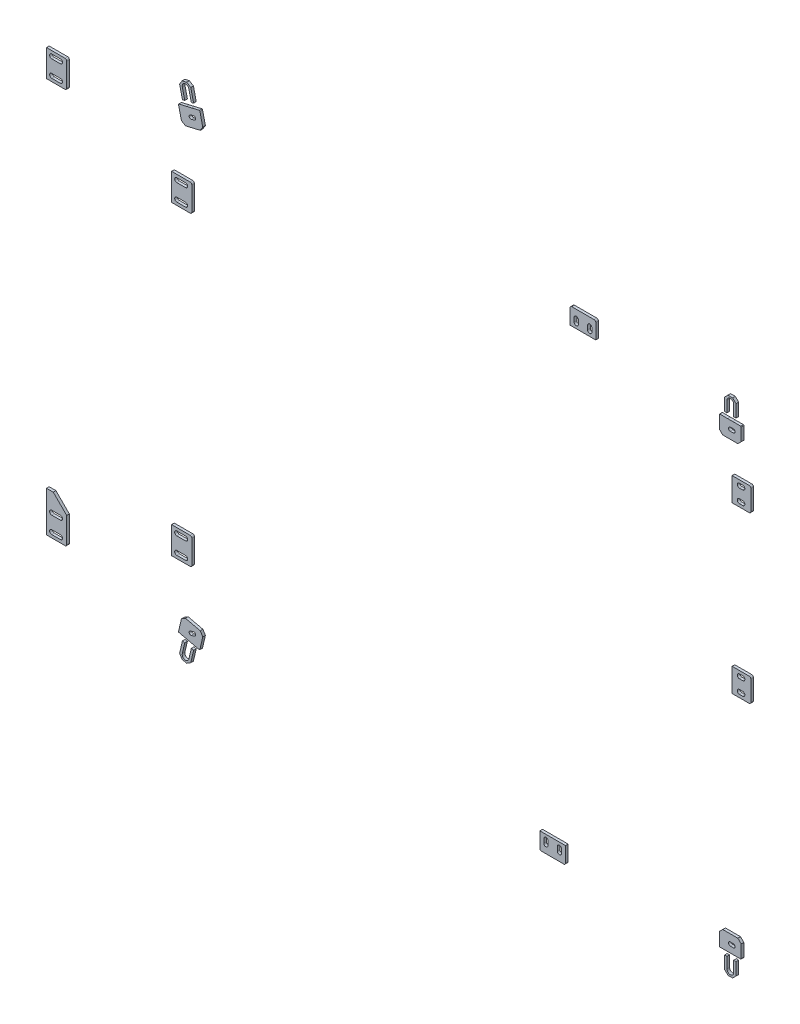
SolidWorks part; units mm, degrees
ref_plane "Plan de face" through (0, 0, 0) normal (0, 0, 1) x (1, 0, 0)
ref_plane "Plan de dessus" through (0, 0, 0) normal (0, 1, 0) x (1, 0, 0)
ref_plane "Plan de droite" through (0, 0, 0) normal (1, 0, 0) x (0, 0, -1)
sketch "CHAMBER" plane through (0, 0, 0) normal (0, 0, 1) x (1, 0, 0)
  line L0 (5467.6161, 2646.2983) -> (5467.6161, 741.2984)
  line L1 (7884.0547, 739.8009) -> (7884.0547, 723.3009)
  line L2 (7851.0547, 723.3009) -> (7851.0547, 739.8009)
  line L3 (7691.0546, 723.3009) -> (7691.0546, 739.8009)
  line L4 (7804.0545, 739.8009) -> (7804.0545, 723.3009)
  line L5 (7771.0545, 723.3009) -> (7771.0545, 737.801)
  line L6 (7853.9546, 714.831) -> (7853.9546, 716.831)
  line L7 (7854.0695, 716.831) -> (7854.3342, 723.3009)
  line L8 (7693.9545, 714.831) -> (7693.9545, 716.831)
  line L9 (7694.0694, 716.831) -> (7694.3341, 723.3009)
  line L10 (7881.1546, 716.831) -> (7881.1546, 714.831)
  line L11 (7880.775, 723.3009) -> (7881.0399, 716.831)
  line L12 (7774.0693, 716.831) -> (7774.334, 723.3009)
  line L13 (7800.7751, 723.3009) -> (7801.0397, 716.831)
  line L14 (7773.9547, 714.831) -> (7773.9547, 716.831)
  line L15 (7801.1547, 716.831) -> (7801.1547, 714.831)
  line L16 (7721.1545, 716.831) -> (7721.1545, 714.831)
  line L17 (7720.7752, 723.3009) -> (7721.0398, 716.831)
  line L18 (8387.6162, 741.2984) -> (5467.6161, 741.2984)
  line L19 (7802.5546, 739.8009) -> (7802.5546, 737.801)
  line L20 (7767.5546, 739.8009) -> (7767.5546, 737.801)
  line L21 (7802.5546, 737.801) -> (7767.5546, 737.801)
  line L22 (7777.5546, 736.801) -> (7777.5546, 737.801)
  line L23 (7777.5546, 736.801) -> (7792.5547, 736.801)
  line L24 (7792.5547, 736.801) -> (7792.5547, 737.801)
  line L25 (8337.5545, 741.2982) -> (8337.5545, 2646.2983)
  line L26 (7723.3296, 723.3009) -> (7691.0546, 723.3009)
  line L27 (7804.0545, 723.3009) -> (7771.0545, 723.3009)
  line L28 (7884.0547, 723.3009) -> (7851.0547, 723.3009)
  line L29 (7853.9546, 714.831) -> (7881.1546, 714.831)
  line L30 (7876.0546, 705.8309) -> (7876.0546, 714.831)
  line L31 (7859.0546, 705.8309) -> (7876.0546, 705.8309)
  line L32 (7721.1545, 716.831) -> (7693.9545, 716.831)
  line L33 (7693.9545, 714.831) -> (7721.1545, 714.831)
  line L34 (7716.0547, 705.8309) -> (7716.0547, 714.831)
  line L35 (7699.0545, 705.8309) -> (7716.0547, 705.8309)
  line L36 (7881.1546, 716.831) -> (7853.9546, 716.831)
  line L37 (7859.0546, 705.8309) -> (7859.0546, 714.831)
  line L38 (7801.1547, 714.831) -> (7773.9547, 714.831)
  line L39 (7773.9547, 716.831) -> (7801.1547, 716.831)
  line L40 (7796.0546, 705.8309) -> (7796.0546, 714.831)
  line L41 (7779.0547, 705.8309) -> (7796.0546, 705.8309)
  line L42 (7779.0547, 705.8309) -> (7779.0547, 714.831)
  line L43 (7699.0545, 705.8309) -> (7699.0545, 714.831)
  line L44 (7724.0544, 739.8009) -> (7724.0544, 723.3009)
  line L45 (6505.8003, 908.756) -> (6734.405, 908.756) construction
  line L46 (7500.2912, 1967.4217) -> (7493.9412, 1967.4217) construction
  line L47 (7493.9412, 1956.3091) -> (7500.2912, 1956.3091) construction
  line L48 (7312.9662, 2506.9748) -> (7417.3912, 2506.9748) construction
  line L49 (7297.0912, 2319.6498) -> (7297.0912, 2548.2498) construction
  line L50 (6505.8003, 2506.9748) -> (6734.405, 2506.9748) construction
  line L51 (6547.08, 2431.0094) -> (6547.08, 2491.0998) construction
  line L52 (6737.58, 2303.7748) -> (6505.782, 2303.7748) construction
  line L53 (6750.28, 2491.0998) -> (6750.28, 2319.6498) construction
  line L54 (7309.7912, 2303.7748) -> (7528.8892, 2303.7748) construction
  line L55 (7528.8662, 2564.1248) -> (7312.9662, 2564.1248) construction
  line L56 (6489.93, 2491.0998) -> (6489.93, 2319.6498) construction
  line L57 (7532.3912, 2451.6848) -> (7532.3912, 2566.6848) construction
  line L58 (7417.3912, 2451.6848) -> (7532.3912, 2451.6848) construction
  line L59 (7300.1392, 2491.0998) -> (7300.1392, 2500.4531) construction
  line L60 (6553.6017, 2503.9268) -> (6562.955, 2503.9268) construction
  line L61 (7309.7912, 2293.818) -> (7316.1412, 2293.818) construction
  line L62 (7316.1412, 2290.3636) -> (7309.7912, 2290.3636) construction
  line L63 (6487.37, 2431.0094) -> (6487.37, 2316.0094) construction
  line L64 (6487.37, 2431.0094) -> (6602.37, 2431.0094) construction
  line L65 (6487.37, 2316.0094) -> (6602.37, 2316.0094) construction
  line L66 (6602.37, 2431.0094) -> (6602.37, 2316.0094) construction
  line L67 (7417.3912, 964.046) -> (7417.3912, 849.046) construction
  line L68 (7532.3912, 964.046) -> (7532.3912, 849.046) construction
  line L69 (7417.3912, 849.046) -> (7532.3912, 849.046) construction
  line L70 (7312.9662, 908.756) -> (7417.3912, 908.756) construction
  line L71 (7528.8662, 851.606) -> (7312.9662, 851.606) construction
  line L72 (7417.3912, 964.046) -> (7532.3912, 964.046) construction
  line L73 (7300.1392, 924.631) -> (7300.1392, 915.2777) construction
  line L74 (7804.1954, 739.8009) -> (7804.1954, 723.3009)
  line L75 (7771.1954, 723.3009) -> (7771.1954, 737.8009)
  line L76 (7851.1956, 723.3009) -> (7851.1956, 739.8009)
  line L77 (7691.1955, 723.3009) -> (7691.1955, 739.8009)
  line L78 (7884.1955, 739.8009) -> (7884.1955, 723.3009)
  line L79 (7694.0954, 714.831) -> (7694.0954, 716.8309)
  line L80 (7721.2953, 716.8309) -> (7721.2953, 714.831)
  line L81 (7694.2103, 716.8309) -> (7694.4749, 723.3009)
  line L82 (7720.916, 723.3009) -> (7721.1807, 716.8309)
  line L83 (7854.0954, 714.831) -> (7854.0954, 716.8309)
  line L84 (7881.2954, 716.8309) -> (7881.2954, 714.831)
  line L85 (7854.2104, 716.8309) -> (7854.475, 723.3009)
  line L86 (7880.9159, 723.3009) -> (7881.1807, 716.8309)
  line L87 (7774.0955, 714.831) -> (7774.0955, 716.8309)
  line L88 (7801.2955, 716.8309) -> (7801.2955, 714.831)
  line L89 (7774.2102, 716.8309) -> (7774.4748, 723.3009)
  line L90 (7800.9159, 723.3009) -> (7801.1806, 716.8309)
  line L91 (5467.6161, 2646.2983) -> (8387.6162, 2646.2983)
  line L92 (7802.6955, 739.8009) -> (7802.6955, 737.8009)
  line L93 (7767.6954, 739.8009) -> (7767.6954, 737.8009)
  line L94 (7802.6955, 737.8009) -> (7767.6954, 737.8009)
  line L95 (7777.6954, 736.801) -> (7777.6954, 737.8009)
  line L96 (7777.6954, 736.801) -> (7792.6955, 736.801)
  line L97 (7792.6955, 736.801) -> (7792.6955, 737.8009)
  line L98 (7723.4704, 723.3009) -> (7691.1955, 723.3009)
  line L99 (7804.1954, 723.3009) -> (7771.1954, 723.3009)
  line L100 (7884.1955, 723.3009) -> (7851.1956, 723.3009)
  line L101 (7854.0954, 714.831) -> (7881.2954, 714.831)
  line L102 (7881.2954, 716.8309) -> (7854.0954, 716.8309)
  line L103 (7859.1954, 705.8309) -> (7876.1954, 705.8309)
  line L104 (7721.2953, 716.8309) -> (7694.0954, 716.8309)
  line L105 (7876.1954, 705.8309) -> (7876.1954, 714.831)
  line L106 (7859.1954, 705.8309) -> (7859.1954, 714.831)
  line L107 (7801.2955, 714.831) -> (7774.0955, 714.831)
  line L108 (7774.0955, 716.8309) -> (7801.2955, 716.8309)
  line L109 (7779.1955, 705.8309) -> (7796.1955, 705.8309)
  line L110 (7796.1955, 705.8309) -> (7796.1955, 714.831)
  line L111 (7779.1955, 705.8309) -> (7779.1955, 714.831)
  line L112 (7694.0954, 714.831) -> (7721.2953, 714.831)
  line L113 (7716.1956, 705.8309) -> (7716.1956, 714.831)
  line L114 (7699.1954, 705.8309) -> (7699.1954, 714.831)
  line L115 (7699.1954, 705.8309) -> (7716.1956, 705.8309)
  line L116 (7724.1952, 739.8009) -> (7724.1952, 723.3009)
  line L117 (7797.3094, 2488.455) -> (7833.2304, 2524.376)
  line L118 (7833.2304, 2488.455) -> (7797.3094, 2524.376)
  line L119 (8244.3494, 2323.355) -> (8280.2704, 2359.276)
  line L120 (8280.2704, 2323.355) -> (8244.3494, 2359.276)
  line L121 (8244.3494, 913.655) -> (8280.2704, 949.576)
  line L122 (8280.2704, 913.655) -> (8244.3494, 949.576)
  line L123 (7797.3094, 913.655) -> (7833.2304, 949.576)
  line L124 (7833.2304, 913.655) -> (7797.3094, 949.576)
  line L125 (8244.3494, 1701.055) -> (8280.2704, 1736.976)
  line L126 (8280.2704, 1701.055) -> (8244.3494, 1736.976)
  line L127 (7462.332, 1491.9653) -> (7487.7321, 1491.9653) construction
  line L128 (7500.432, 1479.2653) -> (7500.432, 1428.4654) construction
  line L129 (7487.7321, 1415.7653) -> (7462.332, 1415.7653) construction
  line L130 (7462.332, 1999.9654) -> (7487.7321, 1999.9654) construction
  line L131 (7500.432, 1987.2653) -> (7500.432, 1936.4653) construction
  line L132 (7487.7321, 1923.7653) -> (7462.332, 1923.7653) construction
  line L133 (6547.2209, 984.7213) -> (6547.2209, 924.6309) construction
  line L134 (6737.7208, 1111.9559) -> (6505.9228, 1111.9559) construction
  line L135 (6750.4208, 924.6309) -> (6750.4208, 1096.0809) construction
  line L136 (7297.2321, 946.8559) -> (6750.4208, 946.8559) construction
  line L137 (7297.2321, 1099.256) -> (6750.4208, 1099.256) construction
  line L138 (7462.332, 2303.7748) -> (7462.332, 1111.9559) construction
  line L139 (7309.9321, 2303.7748) -> (7309.9321, 1111.9559) construction
  line L140 (6737.7208, 2303.7748) -> (6737.7208, 1111.9559) construction
  line L141 (6585.3209, 2303.7748) -> (6585.3209, 1111.9559) construction
  line L142 (6490.0709, 924.6309) -> (6490.0709, 1096.0809) construction
  line L143 (7462.332, 1930.1153) -> (7487.7321, 1930.1153) construction
  line L144 (7494.0821, 1936.4653) -> (7494.0821, 1987.2653) construction
  line L145 (7487.7321, 1993.6153) -> (7462.332, 1993.6153) construction
  line L146 (7462.332, 1422.1153) -> (7487.7321, 1422.1153) construction
  line L147 (7494.0821, 1428.4654) -> (7494.0821, 1479.2653) construction
  line L148 (7487.7321, 1485.6153) -> (7462.332, 1485.6153) construction
  line L149 (7500.432, 1967.4216) -> (7494.0821, 1967.4216) construction
  line L150 (7494.0821, 1956.3091) -> (7500.432, 1956.3091) construction
  line L151 (6487.5108, 984.7213) -> (6487.5108, 1099.7213) construction
  line L152 (6487.5108, 984.7213) -> (6602.5108, 984.7213) construction
  line L153 (6487.5108, 1099.7213) -> (6602.5108, 1099.7213) construction
  line L154 (6602.5108, 984.7213) -> (6602.5108, 1099.7213) construction
  line L155 (7313.107, 2506.9747) -> (7417.5321, 2506.9747) construction
  line L156 (6505.9412, 2506.9747) -> (6734.5459, 2506.9747) construction
  line L157 (6547.2209, 2431.0094) -> (6547.2209, 2491.0998) construction
  line L158 (6737.7208, 2303.7748) -> (6505.9228, 2303.7748) construction
  line L159 (6750.4208, 2491.0998) -> (6750.4208, 2319.6497) construction
  line L160 (7297.2321, 2468.8747) -> (6750.4208, 2468.8747) construction
  line L161 (7297.2321, 2316.4747) -> (6750.4208, 2316.4747) construction
  line L162 (7309.9321, 2303.7748) -> (7529.0301, 2303.7748) construction
  line L163 (6490.0709, 2491.0998) -> (6490.0709, 2319.6497) construction
  line L164 (7544.882, 2319.6497) -> (7544.882, 2548.2498) construction
  line L165 (6553.7426, 2503.9267) -> (6563.0958, 2503.9267) construction
  line L166 (7500.432, 2451.6848) -> (7500.432, 2319.6497) construction
  line L167 (7309.9321, 2293.8179) -> (7316.2821, 2293.8179) construction
  line L168 (7316.2821, 2290.3635) -> (7309.9321, 2290.3635) construction
  line L169 (6487.5108, 2431.0094) -> (6487.5108, 2316.0094) construction
  line L170 (6487.5108, 2431.0094) -> (6602.5108, 2431.0094) construction
  line L171 (6487.5108, 2316.0094) -> (6602.5108, 2316.0094) construction
  line L172 (6602.5108, 2431.0094) -> (6602.5108, 2316.0094) construction
  line L173 (7417.5321, 964.0459) -> (7417.5321, 849.0459) construction
  line L174 (7532.5321, 964.0459) -> (7532.5321, 849.0459) construction
  line L175 (7417.5321, 849.0459) -> (7532.5321, 849.0459) construction
  line L176 (7500.432, 1096.0809) -> (7500.432, 964.0459) construction
  line L177 (7313.107, 908.7559) -> (7417.5321, 908.7559) construction
  line L178 (7309.9321, 1111.9559) -> (7529.0301, 1111.9559) construction
  line L179 (7544.882, 1096.0809) -> (7544.882, 867.4809) construction
  line L180 (7529.007, 851.6059) -> (7313.107, 851.6059) construction
  line L181 (7297.2321, 867.4809) -> (7297.2321, 1096.0809) construction
  line L182 (7417.5321, 964.0459) -> (7532.5321, 964.0459) construction
  line L183 (7300.2801, 924.6309) -> (7300.2801, 915.2776) construction
  line L184 (7417.3912, 2451.6848) -> (7417.3912, 2566.6848) construction
  line L185 (8387.6162, 741.2984) -> (8387.6162, 2646.2983)
  line L186 (8387.6162, 2596.2983) -> (8185.4955, 2596.2983)
  line L187 (7842.8495, 2596.2983) -> (6185.1161, 2596.2983)
  line L188 (8387.6162, 791.2984) -> (8219.4668, 791.2984)
  line L189 (7721.9455, 791.2984) -> (6185.1161, 791.2984)
  line L190 (6185.1161, 2646.2983) -> (6185.1161, 741.2984)
  line L191 (6237.2469, 739.6983) -> (6237.2469, 741.2984) construction
  circle A0 centre (7687.7178, 2505.187) radius 52.524
  arc A1 (6750.28, 1096.081) -> (6734.405, 1111.956) centre (6734.405, 1096.081) ccw construction
  arc A2 (7312.9662, 2506.9748) -> (7297.0912, 2491.0998) centre (7312.9662, 2491.0998) ccw construction
  arc A3 (7297.0912, 2319.6498) -> (7312.9662, 2303.7748) centre (7312.9662, 2319.6498) ccw construction
  arc A4 (6750.28, 2491.0998) -> (6734.405, 2506.9748) centre (6734.405, 2491.0998) ccw construction
  arc A5 (6562.955, 2506.9748) -> (6547.08, 2491.0998) centre (6562.955, 2491.0998) ccw construction
  arc A6 (6547.503, 2316.0094) -> (6562.955, 2303.7748) centre (6562.955, 2319.6498) ccw construction
  arc A7 (6734.405, 2303.7748) -> (6750.28, 2319.6498) centre (6734.405, 2319.6498) ccw construction
  arc A8 (7312.9662, 2564.1248) -> (7297.0912, 2548.2498) centre (7312.9662, 2548.2498) ccw construction
  arc A9 (6489.93, 2319.6498) -> (6505.805, 2303.7748) centre (6505.805, 2319.6498) ccw construction
  arc A10 (6505.8003, 2506.9748) -> (6489.93, 2491.0998) centre (6505.805, 2491.0998) ccw construction
  arc A11 (7297.0912, 924.631) -> (7312.9662, 908.756) centre (7312.9662, 924.631) ccw construction
  circle A12 centre (7474.8912, 879.546) radius 14 construction
  arc A13 (7528.8662, 851.606) -> (7544.7412, 867.481) centre (7528.8662, 867.481) ccw construction
  arc A14 (7297.0912, 867.481) -> (7312.9662, 851.606) centre (7312.9662, 867.481) ccw construction
  circle A15 centre (7474.8912, 879.546) radius 7
  circle A16 centre (6517.87, 1042.106) radius 7
  circle A17 centre (6517.87, 2373.6248) radius 8 construction
  circle A18 centre (7474.8912, 2536.1848) radius 8 construction
  circle A19 centre (8151.1547, 930.387) radius 52.524
  circle A20 centre (7687.8587, 930.387) radius 52.524
  arc A21 (7500.432, 1479.2653) -> (7487.7321, 1491.9653) centre (7487.732, 1479.2653) ccw construction
  arc A22 (7487.7321, 1415.7653) -> (7500.432, 1428.4654) centre (7487.732, 1428.4653) ccw construction
  arc A23 (7500.432, 1987.2653) -> (7487.7321, 1999.9654) centre (7487.732, 1987.2654) ccw construction
  arc A24 (7487.7321, 1923.7653) -> (7500.432, 1936.4653) centre (7487.732, 1936.4653) ccw construction
  arc A25 (6734.5459, 908.7559) -> (6750.4208, 924.6309) centre (6734.5458, 924.6309) ccw construction
  arc A26 (6547.2209, 924.6309) -> (6563.0959, 908.7559) centre (6563.0959, 924.6309) ccw construction
  arc A27 (6563.0959, 1111.9559) -> (6547.6439, 1099.7213) centre (6563.0959, 1096.0809) ccw construction
  arc A28 (6750.4208, 1096.0809) -> (6734.5459, 1111.9559) centre (6734.5458, 1096.0809) ccw construction
  arc A29 (6505.9459, 1111.9559) -> (6490.0709, 1096.0809) centre (6505.9459, 1096.0809) ccw construction
  arc A30 (6490.0709, 924.6309) -> (6505.9459, 908.7559) centre (6505.9459, 924.6309) ccw construction
  arc A31 (7487.7321, 1930.1153) -> (7494.0821, 1936.4653) centre (7487.7321, 1936.4653) ccw construction
  arc A32 (7494.0821, 1987.2653) -> (7487.7321, 1993.6153) centre (7487.7321, 1987.2653) ccw construction
  arc A33 (7487.7321, 1422.1153) -> (7494.0821, 1428.4654) centre (7487.7321, 1428.4653) ccw construction
  arc A34 (7494.0821, 1479.2653) -> (7487.7321, 1485.6153) centre (7487.7321, 1479.2653) ccw construction
  arc A35 (6750.4208, 2491.0998) -> (6734.5459, 2506.9747) centre (6734.5458, 2491.0997) ccw construction
  arc A36 (6563.0959, 2506.9747) -> (6547.2209, 2491.0998) centre (6563.0959, 2491.0997) ccw construction
  arc A37 (6547.6439, 2316.0094) -> (6563.0959, 2303.7747) centre (6563.0959, 2319.6497) ccw construction
  arc A38 (6734.5459, 2303.7747) -> (6750.4208, 2319.6497) centre (6734.5458, 2319.6497) ccw construction
  arc A39 (7544.882, 2548.2498) -> (7529.0071, 2564.1247) centre (7529.007, 2548.2497) ccw construction
  arc A40 (6490.0709, 2319.6497) -> (6505.9459, 2303.7747) centre (6505.9459, 2319.6497) ccw construction
  arc A41 (6505.9412, 2506.9747) -> (6490.0709, 2491.0998) centre (6505.9459, 2491.0997) ccw construction
  arc A42 (7529.0071, 2303.7747) -> (7544.882, 2319.6497) centre (7529.007, 2319.6497) ccw construction
  arc A43 (7484.5571, 2303.7747) -> (7500.432, 2319.6497) centre (7484.557, 2319.6497) ccw construction
  arc A44 (7297.2321, 924.6309) -> (7313.107, 908.7559) centre (7313.1071, 924.6309) ccw construction
  arc A45 (7313.1071, 1111.9559) -> (7297.2321, 1096.0809) centre (7313.1071, 1096.0809) ccw construction
  arc A46 (7529.007, 851.6059) -> (7544.882, 867.4809) centre (7529.007, 867.4809) ccw construction
  arc A47 (7297.2321, 867.4809) -> (7313.107, 851.6059) centre (7313.1071, 867.4809) ccw construction
  arc A48 (7544.882, 1096.0809) -> (7529.0071, 1111.9559) centre (7529.007, 1096.0809) ccw construction
  arc A49 (7500.432, 1096.0809) -> (7484.5571, 1111.9559) centre (7484.557, 1096.0809) ccw construction
  circle A50 centre (8150.6401, 2505.187) radius 52.524
  circle A51 centre (6260.1161, 2621.2983) radius 18.8884
  circle A52 centre (7632.6161, 2621.2983) radius 18.8884
  circle A53 centre (7682.6161, 2621.2983) radius 18.8884
  circle A54 centre (8312.6161, 2621.2983) radius 18.8884
  circle A55 centre (8362.6161, 2621.2984) radius 18.8884
  circle A56 centre (8362.6161, 766.2983) radius 18.8884
  circle A57 centre (8312.6161, 766.2983) radius 18.8884
  circle A58 centre (7682.6161, 766.2983) radius 18.8884
  circle A59 centre (7632.6161, 766.2983) radius 18.8884
  circle A60 centre (6260.1161, 766.2983) radius 18.8884
  text T0 "C" font "ROMANS" height 45.0233
  text T1 "C" font "ROMANS" height 45.0233
  text T2 "C" font "ROMANS" height 45.0233
  text T3 "C" font "ROMANS" height 45.0233
sketch "DATUM" plane through (0, 0, 0) normal (0, 0, 1) x (1, 0, 0)
  line L0 (6538.3155, 1099.8161) -> (6487.5151, 1049.0219)
  line L1 (6487.5151, 1049.0219) -> (6487.5151, 1099.8161)
  line L2 (6487.5151, 1099.8161) -> (6538.3155, 1099.8161)
  line L3 (6538.3113, 2316.0094) -> (6487.5108, 2366.8036)
  line L4 (6487.5108, 2366.8036) -> (6487.5108, 2316.0094)
  line L5 (6487.5108, 2316.0094) -> (6538.3113, 2316.0094)
  line L6 (7481.7316, 2566.6848) -> (7532.5321, 2515.8905)
  line L7 (7532.5321, 2515.8905) -> (7532.5321, 2566.6848)
  line L8 (7532.5321, 2566.6848) -> (7481.7316, 2566.6848)
  line L9 (7481.7316, 848.0323) -> (7532.5321, 898.8265)
  line L10 (7532.5321, 898.8265) -> (7532.5321, 848.0323)
  line L11 (7532.5321, 848.0323) -> (7481.7316, 848.0323)
  line L12 (6185.1161, 791.2984) -> (6235.9103, 741.2984)
  line L13 (6235.9103, 741.2984) -> (6185.1161, 741.2984)
  line L14 (6185.1161, 741.2984) -> (6185.1161, 791.2984)
  line L15 (6185.1161, 2596.2983) -> (6235.9104, 2646.2983)
  line L16 (6235.9104, 2646.2983) -> (6185.1161, 2646.2983)
  line L17 (6185.1161, 2646.2983) -> (6185.1161, 2596.2983)
  circle A0 centre (5467.6161, 2646.2983) radius 38.1
sketch "FLOOR" plane through (0, 0, 0) normal (0, 0, 1) x (1, 0, 0)
  line L0 (7721.9455, 786.8614) -> (8219.4668, 786.8614) construction
  line L1 (8219.4668, 786.8614) -> (8219.4668, 877.26) construction
  line L2 (8219.4668, 877.26) -> (7721.9455, 877.26) construction
  line L3 (7842.8495, 2546.4718) -> (8185.4955, 2546.4718) construction
  line L4 (7890.2537, 1415.4143) -> (7890.2537, 1263.0143) construction
  line L5 (8042.6793, 1263.0143) -> (8042.6539, 1415.4143) construction
  line L6 (8042.6539, 1415.4143) -> (7890.2537, 1415.4143) construction
  line L7 (8042.6793, 1263.0143) -> (7890.2537, 1263.0143) construction
  line L8 (7721.9455, 877.26) -> (7721.9455, 786.8614) construction
  line L9 (7842.8495, 2627.8533) -> (7842.8495, 2546.4718) construction
  line L10 (8185.4955, 2546.4718) -> (8185.4955, 2627.8533) construction
  line L11 (8185.4955, 2627.8533) -> (7842.8495, 2627.8533) construction
  circle A0 centre (6517.87, 2373.6248) radius 14 construction
  circle A1 centre (6517.87, 1042.106) radius 14 construction
  circle A2 centre (7474.8912, 2536.1848) radius 14 construction
  circle A3 centre (7474.8912, 879.546) radius 14 construction
sketch "FRAME-RACK" plane through (0, 0, 0) normal (0, 0, 1) x (1, 0, 0)
  line L0 (7551.0955, 904.987) -> (7641.7438, 904.987) construction
  line L1 (8196.9878, 904.987) -> (8287.6658, 904.987) construction
  line L2 (7843.6239, 2530.587) -> (8105.0398, 2530.587) construction
  line L3 (7551.0955, 2520.7602) -> (7551.0955, 904.987) construction
  line L4 (7551.2363, 904.987) -> (7641.8847, 904.987) construction
  line L5 (7843.7647, 904.987) -> (8105.1807, 904.987) construction
  line L6 (8197.1286, 904.987) -> (8287.8067, 904.987) construction
  line L7 (7551.2363, 2520.7601) -> (7637.6965, 2520.7601) construction
  line L8 (7733.9081, 2530.587) -> (7787.0441, 2530.587) construction
  line L9 (8197.1286, 2530.587) -> (8287.8067, 2530.587) construction
  line L10 (8287.8067, 2530.587) -> (8287.8067, 2368.4851) construction
  line L11 (8287.8067, 2311.6889) -> (8287.8067, 904.987) construction
  line L12 (7733.8326, 904.987) -> (7786.9686, 904.987) construction
sketch "FRONTEND" plane through (0, 0, 0) normal (0, 0, 1) x (1, 0, 0)
  circle A0 centre (6146.1161, 2580.8983) radius 31.75
  circle A1 centre (6146.1161, 806.7083) radius 31.75
  circle A2 centre (5533.0161, 786.7033) radius 31.75
  circle A3 centre (6146.1161, 2580.8983) radius 31.75
  circle A4 centre (5533.0161, 2600.8983) radius 31.75
sketch "SEISMIC" plane through (0, 0, 0) normal (0, 0, 1) x (1, 0, 0)
  line L0 (5723.4344, 2490.8677) -> (5736.1344, 2490.8677)
  line L1 (5736.1344, 2490.8677) -> (5736.1344, 2484.5177)
  line L2 (5723.4344, 2484.5177) -> (5723.4344, 2490.8677)
  line L3 (5736.1344, 2484.5177) -> (5736.1344, 2395.6177)
  line L4 (5723.4344, 2484.5177) -> (5723.4344, 2395.6177)
  line L5 (5736.1344, 2389.2677) -> (5723.4344, 2389.2677)
  line L6 (5736.1344, 2395.6177) -> (5736.1344, 2389.2677)
  line L7 (5723.4344, 2389.2677) -> (5723.4344, 2395.6177)
  line L8 (5742.4844, 2389.2677) -> (5736.1344, 2389.2677)
  line L9 (5736.1344, 2490.8677) -> (5742.4844, 2490.8677)
  line L10 (5812.3344, 2484.5177) -> (5812.3344, 2395.6177)
  line L11 (5755.6924, 2400.3802) -> (5788.7124, 2400.3802)
  line L12 (5788.7124, 2416.2552) -> (5755.6924, 2416.2552)
  line L13 (5788.7124, 2479.7552) -> (5755.6924, 2479.7552)
  line L14 (5755.6924, 2463.8802) -> (5788.7124, 2463.8802)
  line L15 (5742.4844, 2389.2677) -> (5805.9844, 2389.2677)
  line L16 (5742.4844, 2490.8677) -> (5805.9844, 2490.8677)
  line L17 (5717.0844, 2471.8177) -> (5742.4844, 2471.8177)
  line L18 (5717.0844, 2440.0677) -> (5742.4844, 2440.0677)
  line L19 (5717.0844, 2408.3177) -> (5742.4844, 2408.3177)
  line L20 (6166.1752, 2322.6689) -> (6194.7502, 2322.6689)
  line L21 (6166.1752, 2316.3189) -> (6166.1752, 2322.6689)
  line L22 (6194.7502, 2221.0689) -> (6166.1752, 2221.0689)
  line L23 (6166.1752, 2221.0689) -> (6166.1752, 2227.4189)
  line L24 (6166.1752, 2227.4189) -> (6166.1752, 2316.3189)
  line L25 (6194.7502, 2322.6689) -> (6207.4502, 2322.6689)
  line L26 (6207.4502, 2322.6689) -> (6207.4502, 2316.3189)
  line L27 (6194.7502, 2316.3189) -> (6194.7502, 2322.6689)
  line L28 (6207.4502, 2316.3189) -> (6207.4502, 2227.4189)
  line L29 (6194.7502, 2316.3189) -> (6194.7502, 2227.4189)
  line L30 (6207.4502, 2221.0689) -> (6194.7502, 2221.0689)
  line L31 (6207.4502, 2227.4189) -> (6207.4502, 2221.0689)
  line L32 (6194.7502, 2221.0689) -> (6194.7502, 2227.4189)
  line L33 (6213.8002, 2221.0689) -> (6207.4502, 2221.0689)
  line L34 (6207.4502, 2322.6689) -> (6213.8002, 2322.6689)
  line L35 (6283.6502, 2316.3189) -> (6283.6502, 2227.4189)
  line L36 (6227.0082, 2232.1814) -> (6260.0282, 2232.1814)
  line L37 (6260.0282, 2248.0564) -> (6227.0082, 2248.0564)
  line L38 (6260.0282, 2311.5564) -> (6227.0082, 2311.5564)
  line L39 (6227.0082, 2295.6814) -> (6260.0282, 2295.6814)
  line L40 (6213.8002, 2221.0689) -> (6277.3002, 2221.0689)
  line L41 (6213.8002, 2322.6689) -> (6277.3002, 2322.6689)
  line L42 (6159.8252, 2303.6189) -> (6213.8002, 2303.6189)
  line L43 (6159.8252, 2271.8689) -> (6213.8002, 2271.8689)
  line L44 (6159.8252, 2240.1189) -> (6213.8002, 2240.1189)
  line L45 (6166.1752, 1169.8391) -> (6194.7502, 1169.8391)
  line L46 (6166.1752, 1163.4891) -> (6166.1752, 1169.8391)
  line L47 (6194.7502, 1068.2391) -> (6166.1752, 1068.2391)
  line L48 (6166.1752, 1068.2391) -> (6166.1752, 1074.5891)
  line L49 (6166.1752, 1074.5891) -> (6166.1752, 1163.4891)
  line L50 (6194.7502, 1169.8391) -> (6207.4502, 1169.8391)
  line L51 (6207.4502, 1169.8391) -> (6207.4502, 1163.4891)
  line L52 (6194.7502, 1163.4891) -> (6194.7502, 1169.8391)
  line L53 (6207.4502, 1163.4891) -> (6207.4502, 1074.5891)
  line L54 (6194.7502, 1163.4891) -> (6194.7502, 1074.5891)
  line L55 (6207.4502, 1068.2391) -> (6194.7502, 1068.2391)
  line L56 (6207.4502, 1074.5891) -> (6207.4502, 1068.2391)
  line L57 (6194.7502, 1068.2391) -> (6194.7502, 1074.5891)
  line L58 (6213.8002, 1068.2391) -> (6207.4502, 1068.2391)
  line L59 (6207.4502, 1169.8391) -> (6213.8002, 1169.8391)
  line L60 (6283.6502, 1163.4891) -> (6283.6502, 1074.5891)
  line L61 (6227.0082, 1079.3516) -> (6260.0282, 1079.3516)
  line L62 (6260.0282, 1095.2266) -> (6227.0082, 1095.2266)
  line L63 (6260.0282, 1158.7266) -> (6227.0082, 1158.7266)
  line L64 (6227.0082, 1142.8516) -> (6260.0282, 1142.8516)
  line L65 (6213.8002, 1068.2391) -> (6277.3002, 1068.2391)
  line L66 (6213.8002, 1169.8391) -> (6277.3002, 1169.8391)
  line L67 (6159.8252, 1150.7891) -> (6213.8002, 1150.7891)
  line L68 (6159.8252, 1119.0391) -> (6213.8002, 1119.0391)
  line L69 (6159.8252, 1087.2891) -> (6213.8002, 1087.2891)
  line L70 (6289.4953, 2545.3078) -> (6278.4168, 2542.4951)
  line L71 (6263.6594, 2562.6522) -> (6263.4462, 2562.6023)
  line L72 (6283.164, 2567.214) -> (6282.9508, 2567.1642)
  line L73 (6283.164, 2567.214) -> (6269.9751, 2623.6042)
  line L74 (6272.4483, 2624.1827) -> (6285.6373, 2567.7925)
  line L75 (6285.6373, 2567.7925) -> (6283.164, 2567.214)
  line L76 (6237.6473, 2622.5645) -> (6252.2824, 2559.9912)
  line L77 (6247.1213, 2637.8231) -> (6237.6473, 2622.5645)
  line L78 (6264.434, 2641.8723) -> (6247.1213, 2637.8231)
  line L79 (6279.6926, 2632.3984) -> (6264.434, 2641.8723)
  line L80 (6260.9729, 2562.0238) -> (6247.7839, 2618.414)
  line L81 (6252.2824, 2559.9912) -> (6260.9729, 2562.0238)
  line L82 (6285.6373, 2567.7925) -> (6294.3277, 2569.8251)
  line L83 (6294.3277, 2569.8251) -> (6279.6926, 2632.3984)
  line L84 (6250.2572, 2618.9924) -> (6263.4462, 2562.6023)
  line L85 (6263.4462, 2562.6023) -> (6260.9729, 2562.0238)
  line L86 (6263.6594, 2562.6522) -> (6251.6806, 2613.8682)
  line L87 (6270.972, 2618.3803) -> (6282.9508, 2567.1642)
  line L88 (6263.6594, 2562.6522) -> (6282.9508, 2567.1642)
  line L89 (6285.424, 2567.7426) -> (6282.9508, 2567.1642)
  line L90 (6263.6594, 2562.6522) -> (6261.1862, 2562.0737)
  line L91 (6310.9809, 2585.0594) -> (6314.0739, 2571.8349)
  line L92 (6301.459, 2571.493) -> (6297.5723, 2588.1106)
  line L93 (6297.5723, 2588.1106) -> (6310.9809, 2585.0594)
  line L94 (6301.459, 2571.493) -> (6311.8466, 2573.9226)
  line L95 (6297.5723, 2588.1106) -> (6281.5374, 2584.3602)
  line L96 (6285.424, 2567.7426) -> (6301.459, 2571.493)
  line L97 (6241.2646, 2574.9409) -> (6245.1512, 2558.3233)
  line L98 (6257.2995, 2578.6912) -> (6241.2646, 2574.9409)
  line L99 (6245.1512, 2558.3233) -> (6261.1862, 2562.0737)
  line L100 (6230.6002, 2566.2593) -> (6233.6932, 2553.0349)
  line L101 (6230.6002, 2566.2593) -> (6241.2646, 2574.9409)
  line L102 (6234.7636, 2555.8938) -> (6245.1512, 2558.3233)
  line L103 (6259.769, 2497.3111) -> (6315.4172, 2510.3265)
  line L104 (6244.5105, 2506.785) -> (6259.769, 2497.3111)
  line L105 (6244.5105, 2506.785) -> (6233.6932, 2553.0349)
  line L106 (6315.4172, 2510.3265) -> (6324.8912, 2525.5851)
  line L107 (6324.8912, 2525.5851) -> (6314.0739, 2571.8349)
  line L108 (6251.6806, 2613.8682) -> (6252.7494, 2614.1182)
  line L109 (6269.9031, 2618.1303) -> (6270.972, 2618.3803)
  line L110 (7709.2718, 2545.9142) -> (7709.2718, 2628.4662) construction
  line L111 (7709.2718, 2558.6145) -> (7805.7942, 2558.6145) construction
  line L112 (7715.622, 2558.6145) -> (7715.622, 2545.9142) construction
  line L113 (7799.444, 2545.9142) -> (7799.444, 2558.6145) construction
  line L114 (7805.7942, 2628.4662) -> (7805.7942, 2545.9142) construction
  line L115 (7709.2718, 2571.3148) -> (7805.7942, 2571.3148) construction
  line L116 (7724.1947, 2604.3356) -> (7724.1947, 2589.0952) construction
  line L117 (7740.0701, 2589.0952) -> (7740.0701, 2604.3356) construction
  line L118 (7715.622, 2634.8163) -> (7799.444, 2634.8163) construction
  line L119 (7774.9959, 2604.3356) -> (7774.9959, 2589.0952) construction
  line L120 (7790.8713, 2589.0952) -> (7790.8713, 2604.3356) construction
  line L121 (7709.2718, 2545.9142) -> (7805.7942, 2545.9142) construction
  line L122 (8323.9171, 2540.6139) -> (8312.4891, 2540.3981)
  line L123 (8324.1711, 2527.1543) -> (8312.7432, 2526.9385)
  line L124 (8302.7101, 2563.3863) -> (8302.4911, 2563.3863)
  line L125 (8322.7411, 2563.3863) -> (8322.5221, 2563.3863)
  line L126 (8322.7411, 2563.3863) -> (8322.7411, 2621.2983)
  line L127 (8325.2811, 2621.2983) -> (8325.2811, 2563.3863)
  line L128 (8325.2811, 2563.3863) -> (8322.7411, 2563.3863)
  line L129 (8291.0261, 2627.6483) -> (8291.0261, 2563.3863)
  line L130 (8303.7261, 2640.3483) -> (8291.0261, 2627.6483)
  line L131 (8321.5061, 2640.3483) -> (8303.7261, 2640.3483)
  line L132 (8334.2061, 2627.6483) -> (8321.5061, 2640.3483)
  line L133 (8299.9511, 2563.3863) -> (8299.9511, 2621.2983)
  line L134 (8291.0261, 2563.3863) -> (8299.9511, 2563.3863)
  line L135 (8325.2811, 2563.3863) -> (8334.2061, 2563.3863)
  line L136 (8334.2061, 2563.3863) -> (8334.2061, 2627.6483)
  line L137 (8302.4911, 2621.2983) -> (8302.4911, 2563.3863)
  line L138 (8302.4911, 2563.3863) -> (8299.9511, 2563.3863)
  line L139 (8302.7101, 2563.3863) -> (8302.7101, 2615.9846)
  line L140 (8302.7101, 2615.9846) -> (8303.8078, 2615.9846)
  line L141 (8321.4245, 2615.9846) -> (8322.5221, 2615.9846)
  line L142 (8322.5221, 2615.9846) -> (8322.5221, 2563.3863)
  line L143 (8302.7101, 2563.3863) -> (8322.5221, 2563.3863)
  line L144 (8325.0621, 2563.3863) -> (8322.5221, 2563.3863)
  line L145 (8302.7101, 2563.3863) -> (8300.1701, 2563.3863)
  line L146 (8353.8911, 2574.4277) -> (8353.8911, 2560.8463)
  line L147 (8341.5298, 2563.3863) -> (8341.5298, 2580.4524)
  line L148 (8341.5298, 2580.4524) -> (8353.8911, 2574.4277)
  line L149 (8341.5298, 2563.3863) -> (8352.1978, 2563.3863)
  line L150 (8341.5298, 2580.4524) -> (8325.0621, 2580.4524)
  line L151 (8325.0621, 2563.3863) -> (8341.5298, 2563.3863)
  line L152 (8283.7025, 2580.4524) -> (8283.7025, 2563.3863)
  line L153 (8300.1701, 2580.4524) -> (8283.7025, 2580.4524)
  line L154 (8283.7025, 2563.3863) -> (8300.1701, 2563.3863)
  line L155 (8271.3411, 2574.4277) -> (8271.3411, 2560.8463)
  line L156 (8271.3411, 2574.4277) -> (8283.7025, 2580.4524)
  line L157 (8273.0345, 2563.3863) -> (8283.7025, 2563.3863)
  line L158 (8284.0411, 2500.6483) -> (8341.1911, 2500.6483)
  line L159 (8271.3411, 2513.3483) -> (8284.0411, 2500.6483)
  line L160 (8271.3411, 2513.3483) -> (8271.3411, 2560.8463)
  line L161 (8341.1911, 2500.6483) -> (8353.8911, 2513.3483)
  line L162 (8353.8911, 2513.3483) -> (8353.8911, 2560.8463)
  line L163 (8303.6765, 2385.7655) -> (8383.6865, 2385.7655) construction
  line L164 (8383.6865, 2296.8655) -> (8303.6765, 2296.8655) construction
  line L165 (8319.5515, 2385.7655) -> (8319.5515, 2296.8655) construction
  line L166 (8303.6765, 2296.8655) -> (8303.6765, 2385.7655) construction
  line L167 (8359.5565, 2374.653) -> (8346.8565, 2374.653) construction
  line L168 (8346.8565, 2358.778) -> (8359.5565, 2358.778) construction
  line L169 (8390.0365, 2379.4155) -> (8390.0365, 2303.2155) construction
  line L170 (8359.5565, 2323.853) -> (8346.8565, 2323.853) construction
  line L171 (8346.8565, 2307.978) -> (8359.5565, 2307.978) construction
  line L172 (8303.6765, 1763.4655) -> (8383.6865, 1763.4655) construction
  line L173 (8383.6865, 1674.5655) -> (8303.6765, 1674.5655) construction
  line L174 (8319.5515, 1763.4655) -> (8319.5515, 1674.5655) construction
  line L175 (8303.6765, 1674.5655) -> (8303.6765, 1763.4655) construction
  line L176 (8359.5565, 1752.353) -> (8346.8565, 1752.353) construction
  line L177 (8346.8565, 1736.478) -> (8359.5565, 1736.478) construction
  line L178 (8390.0365, 1757.1155) -> (8390.0365, 1680.9155) construction
  line L179 (8359.5565, 1701.553) -> (8346.8565, 1701.553) construction
  line L180 (8346.8565, 1685.678) -> (8359.5565, 1685.678) construction
  line L181 (8323.9171, 846.9828) -> (8312.4891, 847.1985)
  line L182 (8324.1711, 860.4424) -> (8312.7432, 860.6581)
  line L183 (8302.7101, 824.2103) -> (8302.4911, 824.2103)
  line L184 (8322.7411, 824.2103) -> (8322.5221, 824.2103)
  line L185 (8322.7411, 824.2103) -> (8322.7411, 766.2983)
  line L186 (8325.2811, 766.2983) -> (8325.2811, 824.2103)
  line L187 (8325.2811, 824.2103) -> (8322.7411, 824.2103)
  line L188 (8291.0261, 759.9483) -> (8291.0261, 824.2103)
  line L189 (8303.7261, 747.2483) -> (8291.0261, 759.9483)
  line L190 (8321.5061, 747.2483) -> (8303.7261, 747.2483)
  line L191 (8334.2061, 759.9483) -> (8321.5061, 747.2483)
  line L192 (8299.9511, 824.2103) -> (8299.9511, 766.2983)
  line L193 (8291.0261, 824.2103) -> (8299.9511, 824.2103)
  line L194 (8325.2811, 824.2103) -> (8334.2061, 824.2103)
  line L195 (8334.2061, 824.2103) -> (8334.2061, 759.9483)
  line L196 (8302.4911, 766.2983) -> (8302.4911, 824.2103)
  line L197 (8302.4911, 824.2103) -> (8299.9511, 824.2103)
  line L198 (8302.7101, 824.2103) -> (8302.7101, 771.6121)
  line L199 (8302.7101, 771.6121) -> (8303.8078, 771.6121)
  line L200 (8321.4245, 771.6121) -> (8322.5221, 771.6121)
  line L201 (8322.5221, 771.6121) -> (8322.5221, 824.2103)
  line L202 (8302.7101, 824.2103) -> (8322.5221, 824.2103)
  line L203 (8325.0621, 824.2103) -> (8322.5221, 824.2103)
  line L204 (8302.7101, 824.2103) -> (8300.1701, 824.2103)
  line L205 (8353.8911, 813.169) -> (8353.8911, 826.7503)
  line L206 (8341.5298, 824.2103) -> (8341.5298, 807.1443)
  line L207 (8341.5298, 807.1443) -> (8353.8911, 813.169)
  line L208 (8341.5298, 824.2103) -> (8352.1978, 824.2103)
  line L209 (8341.5298, 807.1443) -> (8325.0621, 807.1443)
  line L210 (8325.0621, 824.2103) -> (8341.5298, 824.2103)
  line L211 (8283.7025, 807.1443) -> (8283.7025, 824.2103)
  line L212 (8300.1701, 807.1443) -> (8283.7025, 807.1443)
  line L213 (8283.7025, 824.2103) -> (8300.1701, 824.2103)
  line L214 (8271.3411, 813.169) -> (8271.3411, 826.7503)
  line L215 (8271.3411, 813.169) -> (8283.7025, 807.1443)
  line L216 (8273.0345, 824.2103) -> (8283.7025, 824.2103)
  line L217 (8284.0411, 886.9483) -> (8341.1911, 886.9483)
  line L218 (8271.3411, 874.2483) -> (8284.0411, 886.9483)
  line L219 (8271.3411, 874.2483) -> (8271.3411, 826.7503)
  line L220 (8341.1911, 886.9483) -> (8353.8911, 874.2483)
  line L221 (8353.8911, 874.2483) -> (8353.8911, 826.7503)
  line L222 (5723.4344, 1052.7197) -> (5736.1344, 1052.7197)
  line L223 (5736.1344, 1052.7197) -> (5736.1344, 1046.3697)
  line L224 (5723.4344, 1046.3697) -> (5723.4344, 1052.7197)
  line L225 (5723.4344, 951.1197) -> (5736.1344, 951.1197)
  line L226 (5736.1344, 1046.3697) -> (5736.1344, 951.1197)
  line L227 (5723.4344, 1046.3697) -> (5723.4344, 951.1197)
  line L228 (5736.1344, 900.3197) -> (5723.4344, 900.3197)
  line L229 (5736.1344, 951.1197) -> (5736.1344, 900.3197)
  line L230 (5723.4344, 900.3197) -> (5723.4344, 951.1197)
  line L231 (5742.4844, 900.3197) -> (5736.1344, 900.3197)
  line L232 (5736.1344, 1052.7197) -> (5742.4844, 1052.7197)
  line L233 (5812.3344, 1001.9197) -> (5761.5344, 1052.7197)
  line L234 (5812.3344, 1001.9197) -> (5812.3344, 906.6697)
  line L235 (5755.6924, 911.4322) -> (5788.7124, 911.4322)
  line L236 (5788.7124, 927.3072) -> (5755.6924, 927.3072)
  line L237 (5788.7124, 990.8072) -> (5755.6924, 990.8072)
  line L238 (5755.6924, 974.9322) -> (5788.7124, 974.9322)
  line L239 (5742.4844, 900.3197) -> (5805.9844, 900.3197)
  line L240 (5742.4844, 1052.7197) -> (5761.5344, 1052.7197)
  line L241 (5717.0844, 1033.6697) -> (5742.4844, 1033.6697)
  line L242 (5717.0844, 1001.9197) -> (5742.4844, 1001.9197)
  line L243 (5717.0844, 970.1697) -> (5742.4844, 970.1697)
  line L244 (7601.3729, 889.7858) -> (7601.3729, 877.0855) construction
  line L245 (7691.545, 877.0855) -> (7595.0227, 877.0855) construction
  line L246 (7595.0227, 889.7858) -> (7691.545, 889.7858) construction
  line L247 (7685.1949, 877.0855) -> (7685.1949, 889.7858) construction
  line L248 (7691.545, 864.3852) -> (7595.0227, 864.3852) construction
  line L249 (7691.545, 889.7858) -> (7691.545, 864.3852) construction
  line L250 (7676.6222, 831.3644) -> (7676.6222, 846.6048) construction
  line L251 (7660.7468, 846.6048) -> (7660.7468, 831.3644) construction
  line L252 (7685.1949, 800.8837) -> (7601.3729, 800.8837) construction
  line L253 (7625.821, 831.3644) -> (7625.821, 846.6048) construction
  line L254 (7609.9455, 846.6048) -> (7609.9455, 831.3644) construction
  line L255 (7595.0227, 889.7858) -> (7595.0227, 807.2338) construction
  line L256 (7691.545, 864.3852) -> (7691.545, 807.2338) construction
  line L257 (6292.9464, 848.4273) -> (6281.9895, 845.1731)
  line L258 (6289.1137, 861.3322) -> (6278.1568, 858.078)
  line L259 (6263.6594, 824.9445) -> (6263.4462, 824.9944)
  line L260 (6283.164, 820.3826) -> (6282.9508, 820.4325)
  line L261 (6283.164, 820.3826) -> (6269.9751, 763.9924)
  line L262 (6272.4483, 763.414) -> (6285.6373, 819.8041)
  line L263 (6285.6373, 819.8041) -> (6283.164, 820.3826)
  line L264 (6237.6473, 765.0321) -> (6252.2824, 827.6054)
  line L265 (6247.1213, 749.7736) -> (6237.6473, 765.0321)
  line L266 (6264.434, 745.7243) -> (6247.1213, 749.7736)
  line L267 (6279.6926, 755.1983) -> (6264.434, 745.7243)
  line L268 (6260.9729, 825.5728) -> (6247.7839, 769.1827)
  line L269 (6252.2824, 827.6054) -> (6260.9729, 825.5728)
  line L270 (6285.6373, 819.8041) -> (6294.3277, 817.7716)
  line L271 (6294.3277, 817.7716) -> (6279.6926, 755.1983)
  line L272 (6250.2572, 768.6042) -> (6263.4462, 824.9944)
  line L273 (6263.4462, 824.9944) -> (6260.9729, 825.5728)
  line L274 (6263.6594, 824.9445) -> (6251.6806, 773.7284)
  line L275 (6251.6806, 773.7284) -> (6252.7494, 773.4784)
  line L276 (6269.9031, 769.4664) -> (6270.972, 769.2164)
  line L277 (6270.972, 769.2164) -> (6282.9508, 820.4325)
  line L278 (6263.6594, 824.9445) -> (6282.9508, 820.4325)
  line L279 (6285.424, 819.854) -> (6282.9508, 820.4325)
  line L280 (6263.6594, 824.9445) -> (6261.1862, 825.523)
  line L281 (6310.9809, 802.5372) -> (6314.0739, 815.7617)
  line L282 (6301.459, 816.1037) -> (6297.5723, 799.4861)
  line L283 (6297.5723, 799.4861) -> (6310.9809, 802.5372)
  line L284 (6301.459, 816.1037) -> (6311.8466, 813.6741)
  line L285 (6297.5723, 799.4861) -> (6281.5374, 803.2365)
  line L286 (6285.424, 819.854) -> (6301.459, 816.1037)
  line L287 (6241.2646, 812.6558) -> (6245.1512, 829.2733)
  line L288 (6257.2995, 808.9054) -> (6241.2646, 812.6558)
  line L289 (6245.1512, 829.2733) -> (6261.1862, 825.523)
  line L290 (6230.6002, 821.3373) -> (6233.6932, 834.5618)
  line L291 (6230.6002, 821.3373) -> (6241.2646, 812.6558)
  line L292 (6234.7636, 831.7029) -> (6245.1512, 829.2733)
  line L293 (6259.769, 890.2856) -> (6315.4172, 877.2701)
  line L294 (6244.5105, 880.8116) -> (6259.769, 890.2856)
  line L295 (6244.5105, 880.8116) -> (6233.6932, 834.5618)
  line L296 (6315.4172, 877.2701) -> (6324.8912, 862.0115)
  line L297 (6324.8912, 862.0115) -> (6314.0739, 815.7617)
  arc A0 (5812.3344, 2484.5177) -> (5805.9844, 2490.8677) centre (5805.9844, 2484.5177) ccw
  arc A1 (5805.9844, 2389.2677) -> (5812.3344, 2395.6177) centre (5805.9844, 2395.6177) ccw
  arc A2 (5755.6924, 2416.2552) -> (5755.6924, 2400.3802) centre (5755.6924, 2408.3177) ccw
  arc A3 (5788.7124, 2400.3802) -> (5788.7124, 2416.2552) centre (5788.7124, 2408.3177) ccw
  arc A4 (5788.7124, 2463.8802) -> (5788.7124, 2479.7552) centre (5788.7124, 2471.8177) ccw
  arc A5 (5755.6924, 2479.7552) -> (5755.6924, 2463.8802) centre (5755.6924, 2471.8177) ccw
  arc A6 (6283.6502, 2316.3189) -> (6277.3002, 2322.6689) centre (6277.3002, 2316.3189) ccw
  arc A7 (6277.3002, 2221.0689) -> (6283.6502, 2227.4189) centre (6277.3002, 2227.4189) ccw
  arc A8 (6227.0082, 2248.0564) -> (6227.0082, 2232.1814) centre (6227.0082, 2240.1189) ccw
  arc A9 (6260.0282, 2232.1814) -> (6260.0282, 2248.0564) centre (6260.0282, 2240.1189) ccw
  arc A10 (6260.0282, 2295.6814) -> (6260.0282, 2311.5564) centre (6260.0282, 2303.6189) ccw
  arc A11 (6227.0082, 2311.5564) -> (6227.0082, 2295.6814) centre (6227.0082, 2303.6189) ccw
  arc A12 (6283.6502, 1163.4891) -> (6277.3002, 1169.8391) centre (6277.3002, 1163.4891) ccw
  arc A13 (6277.3002, 1068.2391) -> (6283.6502, 1074.5891) centre (6277.3002, 1074.5891) ccw
  arc A14 (6227.0082, 1095.2266) -> (6227.0082, 1079.3516) centre (6227.0082, 1087.2891) ccw
  arc A15 (6260.0282, 1079.3516) -> (6260.0282, 1095.2266) centre (6260.0282, 1087.2891) ccw
  arc A16 (6260.0282, 1142.8516) -> (6260.0282, 1158.7266) centre (6260.0282, 1150.7891) ccw
  arc A17 (6227.0082, 1158.7266) -> (6227.0082, 1142.8516) centre (6227.0082, 1150.7891) ccw
  circle A18 centre (6280.0731, 2535.9711) radius 25.146
  arc A19 (6292.808, 2532.2598) -> (6289.4953, 2545.3078) centre (6291.1516, 2538.7838) ccw
  arc A20 (6278.4168, 2542.4951) -> (6281.7295, 2529.4471) centre (6280.0731, 2535.9711) ccw
  arc A21 (6272.4483, 2624.1827) -> (6247.7839, 2618.414) centre (6260.1161, 2621.2983) ccw
  arc A22 (6269.9751, 2623.6042) -> (6250.2572, 2618.9924) centre (6260.1161, 2621.2983) ccw
  arc A23 (6252.7494, 2614.1182) -> (6269.9031, 2618.1303) centre (6260.1161, 2621.2983) ccw
  arc A24 (7724.1947, 2589.0952) -> (7740.0701, 2589.0952) centre (7732.1324, 2589.0952) ccw construction
  arc A25 (7740.0701, 2604.3356) -> (7724.1947, 2604.3356) centre (7732.1324, 2604.3356) ccw construction
  arc A26 (7805.7942, 2628.4662) -> (7799.444, 2634.8163) centre (7799.444, 2628.4662) ccw construction
  arc A27 (7715.622, 2634.8163) -> (7709.2718, 2628.4662) centre (7715.622, 2628.4662) ccw construction
  arc A28 (7774.9959, 2589.0952) -> (7790.8713, 2589.0952) centre (7782.9336, 2589.0952) ccw construction
  arc A29 (7790.8713, 2604.3356) -> (7774.9959, 2604.3356) centre (7782.9336, 2604.3356) ccw construction
  circle A30 centre (8312.6161, 2533.6683) radius 25.146
  arc A31 (8324.1711, 2527.1543) -> (8323.9171, 2540.6139) centre (8324.0441, 2533.8841) ccw
  arc A32 (8312.4891, 2540.3981) -> (8312.7432, 2526.9385) centre (8312.6161, 2533.6683) ccw
  arc A33 (8325.2811, 2621.2983) -> (8299.9511, 2621.2983) centre (8312.6161, 2621.2983) ccw
  arc A34 (8322.7411, 2621.2983) -> (8302.4911, 2621.2983) centre (8312.6161, 2621.2983) ccw
  arc A35 (8303.8078, 2615.9846) -> (8321.4245, 2615.9846) centre (8312.6161, 2621.2983) ccw
  arc A36 (8346.8565, 2374.653) -> (8346.8565, 2358.778) centre (8346.8565, 2366.7155) ccw construction
  arc A37 (8359.5565, 2358.778) -> (8359.5565, 2374.653) centre (8359.5565, 2366.7155) ccw construction
  arc A38 (8383.6865, 2296.8655) -> (8390.0365, 2303.2155) centre (8383.6865, 2303.2155) ccw construction
  arc A39 (8390.0365, 2379.4155) -> (8383.6865, 2385.7655) centre (8383.6865, 2379.4155) ccw construction
  arc A40 (8346.8565, 2323.853) -> (8346.8565, 2307.978) centre (8346.8565, 2315.9155) ccw construction
  arc A41 (8359.5565, 2307.978) -> (8359.5565, 2323.853) centre (8359.5565, 2315.9155) ccw construction
  arc A42 (8346.8565, 1752.353) -> (8346.8565, 1736.478) centre (8346.8565, 1744.4155) ccw construction
  arc A43 (8359.5565, 1736.478) -> (8359.5565, 1752.353) centre (8359.5565, 1744.4155) ccw construction
  arc A44 (8383.6865, 1674.5655) -> (8390.0365, 1680.9155) centre (8383.6865, 1680.9155) ccw construction
  arc A45 (8390.0365, 1757.1155) -> (8383.6865, 1763.4655) centre (8383.6865, 1757.1155) ccw construction
  arc A46 (8346.8565, 1701.553) -> (8346.8565, 1685.678) centre (8346.8565, 1693.6155) ccw construction
  arc A47 (8359.5565, 1685.678) -> (8359.5565, 1701.553) centre (8359.5565, 1693.6155) ccw construction
  circle A48 centre (8312.6161, 853.9283) radius 25.146
  arc A49 (8323.9171, 846.9828) -> (8324.1711, 860.4424) centre (8324.0441, 853.7126) ccw
  arc A50 (8312.7432, 860.6581) -> (8312.4891, 847.1985) centre (8312.6161, 853.9283) ccw
  arc A51 (8299.9511, 766.2983) -> (8325.2811, 766.2983) centre (8312.6161, 766.2983) ccw
  arc A52 (8302.4911, 766.2983) -> (8322.7411, 766.2983) centre (8312.6161, 766.2983) ccw
  arc A53 (8321.4245, 771.6121) -> (8303.8078, 771.6121) centre (8312.6161, 766.2983) ccw
  arc A54 (5805.9844, 900.3197) -> (5812.3344, 906.6697) centre (5805.9844, 906.6697) ccw
  arc A55 (5755.6924, 927.3072) -> (5755.6924, 911.4322) centre (5755.6924, 919.3697) ccw
  arc A56 (5788.7124, 911.4322) -> (5788.7124, 927.3072) centre (5788.7124, 919.3697) ccw
  arc A57 (5788.7124, 974.9322) -> (5788.7124, 990.8072) centre (5788.7124, 982.8697) ccw
  arc A58 (5755.6924, 990.8072) -> (5755.6924, 974.9322) centre (5755.6924, 982.8697) ccw
  arc A59 (7676.6222, 846.6048) -> (7660.7468, 846.6048) centre (7668.6845, 846.6048) ccw construction
  arc A60 (7660.7468, 831.3644) -> (7676.6222, 831.3644) centre (7668.6845, 831.3644) ccw construction
  arc A61 (7595.0227, 807.2338) -> (7601.3729, 800.8837) centre (7601.3728, 807.2338) ccw construction
  arc A62 (7685.1949, 800.8837) -> (7691.545, 807.2338) centre (7685.1949, 807.2338) ccw construction
  arc A63 (7625.821, 846.6048) -> (7609.9455, 846.6048) centre (7617.8833, 846.6048) ccw construction
  arc A64 (7609.9455, 831.3644) -> (7625.821, 831.3644) centre (7617.8833, 831.3644) ccw construction
  circle A65 centre (6280.0731, 851.6256) radius 25.146
  arc A66 (6292.9464, 848.4273) -> (6289.1137, 861.3322) centre (6291.0301, 854.8797) ccw
  arc A67 (6278.1568, 858.078) -> (6281.9895, 845.1731) centre (6280.0731, 851.6256) ccw
  arc A68 (6247.7839, 769.1827) -> (6272.4483, 763.414) centre (6260.1161, 766.2983) ccw
  arc A69 (6250.2572, 768.6042) -> (6269.9751, 763.9924) centre (6260.1161, 766.2983) ccw
  arc A70 (6269.9031, 769.4664) -> (6252.7494, 773.4784) centre (6260.1161, 766.2983) ccw
  ellipse E0 centre (6281.3494, 2585.1638) end of major axis (6283.8227, 2585.7423) minor radius 0.8253 (6278.8762, 2584.5853) -> (6281.5374, 2584.3602) ccw
  ellipse E1 centre (6257.1116, 2579.4949) end of major axis (6259.5848, 2580.0733) minor radius 0.8253 (6257.2995, 2578.6912) -> (6259.5848, 2580.0733) ccw
  ellipse E2 centre (6312.4251, 2571.4493) end of major axis (6313.0035, 2568.976) minor radius 1.6933 (6314.0739, 2571.8349) -> (6311.8466, 2573.9226) ccw
  ellipse E3 centre (6235.342, 2553.4205) end of major axis (6235.9205, 2550.9473) minor radius 1.6933 (6234.7636, 2555.8938) -> (6233.6932, 2553.0349) ccw
  ellipse E4 centre (8325.0621, 2581.2777) end of major axis (8327.6021, 2581.2777) minor radius 0.8253 (8322.5221, 2581.2777) -> (8325.0621, 2580.4524) ccw
  ellipse E5 centre (8300.1701, 2581.2777) end of major axis (8302.7101, 2581.2777) minor radius 0.8253 (8300.1701, 2580.4524) -> (8302.7101, 2581.2777) ccw
  ellipse E6 centre (8352.1978, 2560.8463) end of major axis (8352.1978, 2558.3063) minor radius 1.6933 (8353.8911, 2560.8463) -> (8352.1978, 2563.3863) ccw
  ellipse E7 centre (8273.0345, 2560.8463) end of major axis (8273.0345, 2558.3063) minor radius 1.6933 (8273.0345, 2563.3863) -> (8271.3411, 2560.8463) ccw
  ellipse E8 centre (8325.0621, 806.319) end of major axis (8327.6021, 806.319) minor radius 0.8253 (8325.0621, 807.1443) -> (8322.5221, 806.319) ccw
  ellipse E9 centre (8300.1701, 806.319) end of major axis (8302.7101, 806.319) minor radius 0.8253 (8302.7101, 806.319) -> (8300.1701, 807.1443) ccw
  ellipse E10 centre (8352.1978, 826.7503) end of major axis (8352.1978, 829.2903) minor radius 1.6933 (8352.1978, 824.2103) -> (8353.8911, 826.7503) ccw
  ellipse E11 centre (8273.0345, 826.7503) end of major axis (8273.0345, 829.2903) minor radius 1.6933 (8271.3411, 826.7503) -> (8273.0345, 824.2103) ccw
  ellipse E12 centre (6281.3494, 802.4329) end of major axis (6283.8227, 801.8544) minor radius 0.8253 (6281.5374, 803.2365) -> (6278.8762, 803.0113) ccw
  ellipse E13 centre (6257.1116, 808.1018) end of major axis (6259.5848, 807.5233) minor radius 0.8253 (6259.5848, 807.5233) -> (6257.2995, 808.9054) ccw
  ellipse E14 centre (6312.4251, 816.1474) end of major axis (6313.0035, 818.6206) minor radius 1.6933 (6311.8466, 813.6741) -> (6314.0739, 815.7617) ccw
  ellipse E15 centre (6235.342, 834.1761) end of major axis (6235.9205, 836.6494) minor radius 1.6933 (6233.6932, 834.5618) -> (6234.7636, 831.7029) ccw
sketch "TieDown" plane through (0, 0, 0) normal (0, 0, 1) x (1, 0, 0)
  circle A0 centre (8265.7444, 2547.3045) radius 5.0703
  circle A1 centre (8314.6111, 2533.6401) radius 5.0703
  circle A2 centre (7783.0244, 2596.7105) radius 5.0703
  circle A3 centre (7732.1778, 2596.713) radius 5.0703
  circle A4 centre (6237.541, 2303.6182) radius 5.0703
  circle A5 centre (8314.6249, 853.6872) radius 6 construction
  circle A6 centre (8265.5986, 840.1741) radius 6 construction
  circle A7 centre (7668.7217, 838.9882) radius 5.0703
  circle A8 centre (8314.6249, 853.6872) radius 5.0703
  circle A9 centre (8265.5986, 840.1741) radius 5.0703
  circle A10 centre (6285.5162, 2537.4783) radius 6 construction
  circle A11 centre (6234.7162, 2537.4783) radius 6 construction
  circle A12 centre (6234.7162, 2537.4783) radius 5.0703
  circle A13 centre (6285.5162, 2537.4783) radius 5.0703
  circle A14 centre (5761.418, 982.869) radius 6 construction
  circle A15 centre (5761.418, 982.869) radius 5.0703
  circle A16 centre (5761.418, 919.369) radius 6 construction
  circle A17 centre (5761.418, 919.369) radius 5.0703
  circle A18 centre (6234.8431, 853.2399) radius 6 construction
  circle A19 centre (6234.8431, 853.2399) radius 5.0703
  circle A20 centre (6285.6431, 853.2399) radius 6 construction
  circle A21 centre (6285.6431, 853.2399) radius 5.0703
  circle A22 centre (6237.541, 1087.2884) radius 6 construction
  circle A23 centre (6237.541, 1087.2884) radius 5.0703
  circle A24 centre (6237.541, 1150.7884) radius 6 construction
  circle A25 centre (6237.541, 1150.7884) radius 5.0703
  circle A26 centre (5761.418, 2471.817) radius 5.0703
  circle A27 centre (5761.418, 2408.317) radius 5.0703
  circle A28 centre (6237.541, 2240.1182) radius 5.0703
  circle A29 centre (8353.2065, 1693.6155) radius 6 construction
  circle A30 centre (8353.2065, 2315.9155) radius 6
  circle A31 centre (8353.2065, 2366.7155) radius 6
  circle A32 centre (8353.2065, 1693.6155) radius 5.053 construction
  circle A33 centre (8353.2065, 2366.7155) radius 5.053
  circle A34 centre (8353.2065, 2315.9155) radius 5.053
  circle A35 centre (7617.875, 838.9907) radius 5.0703
  circle A36 centre (8353.2065, 1744.4155) radius 6 construction
  circle A37 centre (8353.2065, 1744.4155) radius 5.053 construction
extrude "Boss.-Extru.1" add sketch "SEISMIC" along normal blind 10
sketch "Esquisse9" plane through (0, 0, 0) normal (0, 0, 1) x (1, 0, 0)
  line L0 (6257.2995, 2578.6912) -> (6241.2646, 2574.9409) construction
  line L1 (6297.5723, 2588.1106) -> (6281.5374, 2584.3602) construction
  line L2 (6310.9809, 2585.0594) -> (6314.0739, 2571.8349) construction
  line L3 (6297.5723, 2588.1106) -> (6310.9809, 2585.0594) construction
  line L4 (6324.8912, 2525.5851) -> (6314.0739, 2571.8349) construction
  line L5 (6315.4172, 2510.3265) -> (6324.8912, 2525.5851) construction
  line L6 (6259.769, 2497.3111) -> (6315.4172, 2510.3265) construction
  line L7 (6244.5105, 2506.785) -> (6259.769, 2497.3111) construction
  line L8 (6244.5105, 2506.785) -> (6233.6932, 2553.0349) construction
  line L9 (6301.459, 2571.493) -> (6311.8466, 2573.9226) construction
  line L10 (8341.5298, 2580.4524) -> (8325.0621, 2580.4524) construction
  line L11 (6230.6002, 2566.2593) -> (6233.6932, 2553.0349) construction
  line L12 (6230.6002, 2566.2593) -> (6241.2646, 2574.9409) construction
  line L13 (6234.7636, 2555.8938) -> (6245.1512, 2558.3233) construction
  line L14 (8300.1701, 2580.4524) -> (8283.7025, 2580.4524) construction
  line L15 (8353.8911, 2574.4277) -> (8353.8911, 2560.8463) construction
  line L16 (8341.5298, 2580.4524) -> (8353.8911, 2574.4277) construction
  line L17 (8353.8911, 2513.3483) -> (8353.8911, 2560.8463) construction
  line L18 (8341.1911, 2500.6483) -> (8353.8911, 2513.3483) construction
  line L19 (8284.0411, 2500.6483) -> (8341.1911, 2500.6483) construction
  line L20 (8271.3411, 2513.3483) -> (8284.0411, 2500.6483) construction
  line L21 (8271.3411, 2513.3483) -> (8271.3411, 2560.8463) construction
  line L22 (8341.5298, 2563.3863) -> (8352.1978, 2563.3863) construction
  line L23 (5717.0844, 2471.8177) -> (5742.4844, 2471.8177) construction
  line L24 (5723.4344, 2490.8677) -> (5736.1344, 2490.8677) construction
  line L25 (5723.4344, 2484.5177) -> (5723.4344, 2490.8677) construction
  line L26 (5723.4344, 2484.5177) -> (5723.4344, 2395.6177) construction
  line L27 (5723.4344, 2389.2677) -> (5723.4344, 2395.6177) construction
  line L28 (5736.1344, 2389.2677) -> (5723.4344, 2389.2677) construction
  line L29 (5736.1344, 2490.8677) -> (5736.1344, 2484.5177) construction
  line L30 (5736.1344, 2484.5177) -> (5736.1344, 2395.6177) construction
  line L31 (5736.1344, 2395.6177) -> (5736.1344, 2389.2677) construction
  line L32 (5742.4844, 2389.2677) -> (5736.1344, 2389.2677) construction
  line L33 (5742.4844, 2389.2677) -> (5805.9844, 2389.2677) construction
  line L34 (5812.3344, 2484.5177) -> (5812.3344, 2395.6177) construction
  line L35 (5742.4844, 2490.8677) -> (5805.9844, 2490.8677) construction
  line L36 (5736.1344, 2490.8677) -> (5742.4844, 2490.8677) construction
  line L37 (8341.5298, 807.1443) -> (8325.0621, 807.1443) construction
  line L38 (8271.3411, 2574.4277) -> (8271.3411, 2560.8463) construction
  line L39 (8271.3411, 2574.4277) -> (8283.7025, 2580.4524) construction
  line L40 (8273.0345, 2563.3863) -> (8283.7025, 2563.3863) construction
  line L41 (6194.7502, 2322.6689) -> (6207.4502, 2322.6689) construction
  line L42 (6207.4502, 2322.6689) -> (6207.4502, 2316.3189) construction
  line L43 (6207.4502, 2316.3189) -> (6207.4502, 2227.4189) construction
  line L44 (6207.4502, 2227.4189) -> (6207.4502, 2221.0689) construction
  line L45 (6213.8002, 2221.0689) -> (6207.4502, 2221.0689) construction
  line L46 (6213.8002, 2221.0689) -> (6277.3002, 2221.0689) construction
  line L47 (6283.6502, 2316.3189) -> (6283.6502, 2227.4189) construction
  line L48 (6213.8002, 2322.6689) -> (6277.3002, 2322.6689) construction
  line L49 (6207.4502, 2322.6689) -> (6213.8002, 2322.6689) construction
  line L50 (6166.1752, 2322.6689) -> (6194.7502, 2322.6689) construction
  line L51 (6166.1752, 2316.3189) -> (6166.1752, 2322.6689) construction
  line L52 (6166.1752, 2227.4189) -> (6166.1752, 2316.3189) construction
  line L53 (6166.1752, 2221.0689) -> (6166.1752, 2227.4189) construction
  line L54 (6194.7502, 2221.0689) -> (6166.1752, 2221.0689) construction
  line L55 (6207.4502, 2221.0689) -> (6194.7502, 2221.0689) construction
  line L56 (6194.7502, 2316.3189) -> (6194.7502, 2322.6689) construction
  line L57 (6194.7502, 2316.3189) -> (6194.7502, 2227.4189) construction
  line L58 (6194.7502, 2221.0689) -> (6194.7502, 2227.4189) construction
  line L59 (5717.0844, 2408.3177) -> (5742.4844, 2408.3177) construction
  line L60 (5717.0844, 2440.0677) -> (5742.4844, 2440.0677) construction
  line L61 (8300.1701, 807.1443) -> (8283.7025, 807.1443) construction
  line L62 (8271.3411, 813.169) -> (8271.3411, 826.7503) construction
  line L63 (8271.3411, 813.169) -> (8283.7025, 807.1443) construction
  line L64 (8353.8911, 874.2483) -> (8353.8911, 826.7503) construction
  line L65 (8341.1911, 886.9483) -> (8353.8911, 874.2483) construction
  line L66 (8284.0411, 886.9483) -> (8341.1911, 886.9483) construction
  line L67 (8271.3411, 874.2483) -> (8284.0411, 886.9483) construction
  line L68 (8271.3411, 874.2483) -> (8271.3411, 826.7503) construction
  line L69 (8273.0345, 824.2103) -> (8283.7025, 824.2103) construction
  line L70 (8353.8911, 813.169) -> (8353.8911, 826.7503) construction
  line L71 (8341.5298, 807.1443) -> (8353.8911, 813.169) construction
  line L72 (8341.5298, 824.2103) -> (8352.1978, 824.2103) construction
  line L73 (6194.7502, 1169.8391) -> (6207.4502, 1169.8391) construction
  line L74 (6207.4502, 1169.8391) -> (6207.4502, 1163.4891) construction
  line L75 (6207.4502, 1163.4891) -> (6207.4502, 1074.5891) construction
  line L76 (6207.4502, 1074.5891) -> (6207.4502, 1068.2391) construction
  line L77 (6213.8002, 1068.2391) -> (6207.4502, 1068.2391) construction
  line L78 (6213.8002, 1068.2391) -> (6277.3002, 1068.2391) construction
  line L79 (6283.6502, 1163.4891) -> (6283.6502, 1074.5891) construction
  line L80 (6213.8002, 1169.8391) -> (6277.3002, 1169.8391) construction
  line L81 (6207.4502, 1169.8391) -> (6213.8002, 1169.8391) construction
  line L82 (6166.1752, 1169.8391) -> (6194.7502, 1169.8391) construction
  line L83 (6166.1752, 1163.4891) -> (6166.1752, 1169.8391) construction
  line L84 (6166.1752, 1074.5891) -> (6166.1752, 1163.4891) construction
  line L85 (6166.1752, 1068.2391) -> (6166.1752, 1074.5891) construction
  line L86 (6194.7502, 1068.2391) -> (6166.1752, 1068.2391) construction
  line L87 (6207.4502, 1068.2391) -> (6194.7502, 1068.2391) construction
  line L88 (6194.7502, 1163.4891) -> (6194.7502, 1169.8391) construction
  line L89 (6194.7502, 1163.4891) -> (6194.7502, 1074.5891) construction
  line L90 (6194.7502, 1068.2391) -> (6194.7502, 1074.5891) construction
  line L91 (6159.8252, 2240.1189) -> (6213.8002, 2240.1189) construction
  line L92 (6159.8252, 2271.8689) -> (6213.8002, 2271.8689) construction
  line L93 (6159.8252, 2303.6189) -> (6213.8002, 2303.6189) construction
  line L94 (6257.2995, 808.9054) -> (6241.2646, 812.6558) construction
  line L95 (6297.5723, 799.4861) -> (6281.5374, 803.2365) construction
  line L96 (6283.164, 2567.214) -> (6282.9508, 2567.1642) construction
  line L97 (6283.164, 2567.214) -> (6269.9751, 2623.6042) construction
  line L98 (6250.2572, 2618.9924) -> (6263.4462, 2562.6023) construction
  line L99 (6285.6373, 2567.7925) -> (6283.164, 2567.214) construction
  line L100 (6263.6594, 2562.6522) -> (6263.4462, 2562.6023) construction
  line L101 (6263.4462, 2562.6023) -> (6260.9729, 2562.0238) construction
  line L102 (6263.6594, 2562.6522) -> (6251.6806, 2613.8682) construction
  line L103 (6251.6806, 2613.8682) -> (6252.7494, 2614.1182) construction
  line L104 (6269.9031, 2618.1303) -> (6270.972, 2618.3803) construction
  line L105 (6270.972, 2618.3803) -> (6282.9508, 2567.1642) construction
  line L106 (6263.6594, 2562.6522) -> (6282.9508, 2567.1642) construction
  line L107 (6263.6594, 2562.6522) -> (6261.1862, 2562.0737) construction
  line L108 (6245.1512, 2558.3233) -> (6261.1862, 2562.0737) construction
  line L109 (6159.8252, 1087.2891) -> (6213.8002, 1087.2891) construction
  line L110 (6159.8252, 1119.0391) -> (6213.8002, 1119.0391) construction
  line L111 (6159.8252, 1150.7891) -> (6213.8002, 1150.7891) construction
  line L112 (6230.6002, 821.3373) -> (6233.6932, 834.5618) construction
  line L113 (6230.6002, 821.3373) -> (6241.2646, 812.6558) construction
  line L114 (6244.5105, 880.8116) -> (6233.6932, 834.5618) construction
  line L115 (6244.5105, 880.8116) -> (6259.769, 890.2856) construction
  line L116 (6259.769, 890.2856) -> (6315.4172, 877.2701) construction
  line L117 (6315.4172, 877.2701) -> (6324.8912, 862.0115) construction
  line L118 (6324.8912, 862.0115) -> (6314.0739, 815.7617) construction
  line L119 (6234.7636, 831.7029) -> (6245.1512, 829.2733) construction
  line L120 (6310.9809, 802.5372) -> (6314.0739, 815.7617) construction
  line L121 (6297.5723, 799.4861) -> (6310.9809, 802.5372) construction
  line L122 (6301.459, 816.1037) -> (6311.8466, 813.6741) construction
  line L123 (6301.459, 2571.493) -> (6297.5723, 2588.1106) construction
  line L124 (6285.424, 2567.7426) -> (6282.9508, 2567.1642) construction
  line L125 (6285.424, 2567.7426) -> (6301.459, 2571.493) construction
  line L126 (6272.4483, 2624.1827) -> (6285.6373, 2567.7925) construction
  line L127 (6260.9729, 2562.0238) -> (6247.7839, 2618.414) construction
  line L128 (6252.2824, 2559.9912) -> (6260.9729, 2562.0238) construction
  line L129 (6237.6473, 2622.5645) -> (6252.2824, 2559.9912) construction
  line L130 (6247.1213, 2637.8231) -> (6237.6473, 2622.5645) construction
  line L131 (6264.434, 2641.8723) -> (6247.1213, 2637.8231) construction
  line L132 (6279.6926, 2632.3984) -> (6264.434, 2641.8723) construction
  line L133 (6294.3277, 2569.8251) -> (6279.6926, 2632.3984) construction
  line L134 (6285.6373, 2567.7925) -> (6294.3277, 2569.8251) construction
  line L135 (6241.2646, 2574.9409) -> (6245.1512, 2558.3233) construction
  line L136 (8325.2811, 2621.2983) -> (8325.2811, 2563.3863) construction
  line L137 (8299.9511, 2563.3863) -> (8299.9511, 2621.2983) construction
  line L138 (8291.0261, 2563.3863) -> (8299.9511, 2563.3863) construction
  line L139 (8291.0261, 2627.6483) -> (8291.0261, 2563.3863) construction
  line L140 (8303.7261, 2640.3483) -> (8291.0261, 2627.6483) construction
  line L141 (8321.5061, 2640.3483) -> (8303.7261, 2640.3483) construction
  line L142 (8334.2061, 2627.6483) -> (8321.5061, 2640.3483) construction
  line L143 (8334.2061, 2563.3863) -> (8334.2061, 2627.6483) construction
  line L144 (8325.2811, 2563.3863) -> (8334.2061, 2563.3863) construction
  line L145 (8302.4911, 2563.3863) -> (8299.9511, 2563.3863) construction
  line L146 (8325.2811, 2563.3863) -> (8322.7411, 2563.3863) construction
  line L147 (8322.7411, 2563.3863) -> (8322.5221, 2563.3863) construction
  line L148 (8302.7101, 2563.3863) -> (8302.7101, 2615.9846) construction
  line L149 (8302.7101, 2615.9846) -> (8303.8078, 2615.9846) construction
  line L150 (8321.4245, 2615.9846) -> (8322.5221, 2615.9846) construction
  line L151 (8322.5221, 2615.9846) -> (8322.5221, 2563.3863) construction
  line L152 (8302.7101, 2563.3863) -> (8322.5221, 2563.3863) construction
  line L153 (8325.0621, 2563.3863) -> (8322.5221, 2563.3863) construction
  line L154 (8325.0621, 2563.3863) -> (8341.5298, 2563.3863) construction
  line L155 (8322.7411, 2563.3863) -> (8322.7411, 2621.2983) construction
  line L156 (8302.4911, 2621.2983) -> (8302.4911, 2563.3863) construction
  line L157 (8302.7101, 2563.3863) -> (8302.4911, 2563.3863) construction
  line L158 (8302.7101, 2563.3863) -> (8300.1701, 2563.3863) construction
  line L159 (8283.7025, 2563.3863) -> (8300.1701, 2563.3863) construction
  line L160 (8283.7025, 2580.4524) -> (8283.7025, 2563.3863) construction
  line L161 (8341.5298, 2563.3863) -> (8341.5298, 2580.4524) construction
  line L162 (6289.4953, 2545.3078) -> (6278.4168, 2542.4951) construction
  line L163 (8325.2811, 766.2983) -> (8325.2811, 824.2103) construction
  line L164 (8299.9511, 824.2103) -> (8299.9511, 766.2983) construction
  line L165 (8291.0261, 824.2103) -> (8299.9511, 824.2103) construction
  line L166 (8291.0261, 759.9483) -> (8291.0261, 824.2103) construction
  line L167 (8303.7261, 747.2483) -> (8291.0261, 759.9483) construction
  line L168 (8321.5061, 747.2483) -> (8303.7261, 747.2483) construction
  line L169 (8334.2061, 759.9483) -> (8321.5061, 747.2483) construction
  line L170 (8334.2061, 824.2103) -> (8334.2061, 759.9483) construction
  line L171 (8325.2811, 824.2103) -> (8334.2061, 824.2103) construction
  line L172 (8302.4911, 824.2103) -> (8299.9511, 824.2103) construction
  line L173 (8325.2811, 824.2103) -> (8322.7411, 824.2103) construction
  line L174 (8322.7411, 824.2103) -> (8322.5221, 824.2103) construction
  line L175 (8302.7101, 824.2103) -> (8302.7101, 771.6121) construction
  line L176 (8302.7101, 771.6121) -> (8303.8078, 771.6121) construction
  line L177 (8321.4245, 771.6121) -> (8322.5221, 771.6121) construction
  line L178 (8322.5221, 771.6121) -> (8322.5221, 824.2103) construction
  line L179 (8302.7101, 824.2103) -> (8322.5221, 824.2103) construction
  line L180 (8325.0621, 824.2103) -> (8322.5221, 824.2103) construction
  line L181 (8325.0621, 824.2103) -> (8341.5298, 824.2103) construction
  line L182 (8322.7411, 824.2103) -> (8322.7411, 766.2983) construction
  line L183 (8302.4911, 766.2983) -> (8302.4911, 824.2103) construction
  line L184 (8302.7101, 824.2103) -> (8302.4911, 824.2103) construction
  line L185 (8302.7101, 824.2103) -> (8300.1701, 824.2103) construction
  line L186 (8283.7025, 824.2103) -> (8300.1701, 824.2103) construction
  line L187 (5723.4344, 1052.7197) -> (5736.1344, 1052.7197) construction
  line L188 (5723.4344, 1046.3697) -> (5723.4344, 1052.7197) construction
  line L189 (5723.4344, 1046.3697) -> (5723.4344, 951.1197) construction
  line L190 (5736.1344, 1052.7197) -> (5736.1344, 1046.3697) construction
  line L191 (5736.1344, 1046.3697) -> (5736.1344, 951.1197) construction
  line L192 (5736.1344, 1052.7197) -> (5742.4844, 1052.7197) construction
  line L193 (5742.4844, 1052.7197) -> (5761.5344, 1052.7197) construction
  line L194 (5812.3344, 1001.9197) -> (5761.5344, 1052.7197) construction
  line L195 (5812.3344, 1001.9197) -> (5812.3344, 906.6697) construction
  line L196 (5742.4844, 900.3197) -> (5805.9844, 900.3197) construction
  line L197 (5742.4844, 900.3197) -> (5736.1344, 900.3197) construction
  line L198 (8283.7025, 807.1443) -> (8283.7025, 824.2103) construction
  line L199 (8341.5298, 824.2103) -> (8341.5298, 807.1443) construction
  line L200 (5717.0844, 970.1697) -> (5742.4844, 970.1697) construction
  line L201 (5717.0844, 1001.9197) -> (5742.4844, 1001.9197) construction
  line L202 (5717.0844, 1033.6697) -> (5742.4844, 1033.6697) construction
  line L203 (5736.1344, 900.3197) -> (5723.4344, 900.3197) construction
  line L204 (5723.4344, 900.3197) -> (5723.4344, 951.1197) construction
  line L205 (5736.1344, 951.1197) -> (5736.1344, 900.3197) construction
  line L206 (5723.4344, 951.1197) -> (5736.1344, 951.1197) construction
  line L207 (6272.4483, 763.414) -> (6285.6373, 819.8041) construction
  line L208 (6260.9729, 825.5728) -> (6247.7839, 769.1827) construction
  line L209 (6285.6373, 819.8041) -> (6283.164, 820.3826) construction
  line L210 (6252.2824, 827.6054) -> (6260.9729, 825.5728) construction
  line L211 (6237.6473, 765.0321) -> (6252.2824, 827.6054) construction
  line L212 (6247.1213, 749.7736) -> (6237.6473, 765.0321) construction
  line L213 (6264.434, 745.7243) -> (6247.1213, 749.7736) construction
  line L214 (6279.6926, 755.1983) -> (6264.434, 745.7243) construction
  line L215 (6294.3277, 817.7716) -> (6279.6926, 755.1983) construction
  line L216 (6285.6373, 819.8041) -> (6294.3277, 817.7716) construction
  line L217 (6283.164, 820.3826) -> (6282.9508, 820.4325) construction
  line L218 (6263.6594, 824.9445) -> (6251.6806, 773.7284) construction
  line L219 (6251.6806, 773.7284) -> (6252.7494, 773.4784) construction
  line L220 (6269.9031, 769.4664) -> (6270.972, 769.2164) construction
  line L221 (6270.972, 769.2164) -> (6282.9508, 820.4325) construction
  line L222 (6263.6594, 824.9445) -> (6282.9508, 820.4325) construction
  line L223 (6285.424, 819.854) -> (6282.9508, 820.4325) construction
  line L224 (6285.424, 819.854) -> (6301.459, 816.1037) construction
  line L225 (6283.164, 820.3826) -> (6269.9751, 763.9924) construction
  line L226 (6250.2572, 768.6042) -> (6263.4462, 824.9944) construction
  line L227 (6263.6594, 824.9445) -> (6263.4462, 824.9944) construction
  line L228 (6263.4462, 824.9944) -> (6260.9729, 825.5728) construction
  line L229 (6263.6594, 824.9445) -> (6261.1862, 825.523) construction
  line L230 (6245.1512, 829.2733) -> (6261.1862, 825.523) construction
  line L231 (6241.2646, 812.6558) -> (6245.1512, 829.2733) construction
  line L232 (6301.459, 816.1037) -> (6297.5723, 799.4861) construction
  line L233 (5788.7124, 990.8072) -> (5755.6924, 990.8072) construction
  line L234 (5755.6924, 974.9322) -> (5788.7124, 974.9322) construction
  line L235 (6292.9464, 848.4273) -> (6281.9895, 845.1731) construction
  line L236 (6289.1137, 861.3322) -> (6278.1568, 858.078) construction
  line L237 (5755.6924, 2400.3802) -> (5788.7124, 2400.3802) construction
  line L238 (5788.7124, 2416.2552) -> (5755.6924, 2416.2552) construction
  line L239 (6227.0082, 2232.1814) -> (6260.0282, 2232.1814) construction
  line L240 (6260.0282, 2248.0564) -> (6227.0082, 2248.0564) construction
  line L241 (5788.7124, 2479.7552) -> (5755.6924, 2479.7552) construction
  line L242 (5755.6924, 2463.8802) -> (5788.7124, 2463.8802) construction
  line L243 (6227.0082, 1079.3516) -> (6260.0282, 1079.3516) construction
  line L244 (6260.0282, 1095.2266) -> (6227.0082, 1095.2266) construction
  line L245 (6260.0282, 2311.5564) -> (6227.0082, 2311.5564) construction
  line L246 (6227.0082, 2295.6814) -> (6260.0282, 2295.6814) construction
  line L247 (6260.0282, 1158.7266) -> (6227.0082, 1158.7266) construction
  line L248 (6227.0082, 1142.8516) -> (6260.0282, 1142.8516) construction
  line L249 (8323.9171, 2540.6139) -> (8312.4891, 2540.3981) construction
  line L250 (8324.1711, 2527.1543) -> (8312.7432, 2526.9385) construction
  line L251 (8323.9171, 846.9828) -> (8312.4891, 847.1985) construction
  line L252 (8324.1711, 860.4424) -> (8312.7432, 860.6581) construction
  line L253 (5755.6924, 911.4322) -> (5788.7124, 911.4322) construction
  line L254 (5788.7124, 927.3072) -> (5755.6924, 927.3072) construction
  line L255 (6257.2995, 2578.6912) -> (6241.2646, 2574.9409)
  line L256 (6297.5723, 2588.1106) -> (6281.5374, 2584.3602)
  line L257 (6310.9809, 2585.0594) -> (6314.0739, 2571.8349)
  line L258 (6297.5723, 2588.1106) -> (6310.9809, 2585.0594)
  line L259 (6324.8912, 2525.5851) -> (6314.0739, 2571.8349)
  line L260 (6315.4172, 2510.3265) -> (6324.8912, 2525.5851)
  line L261 (6259.769, 2497.3111) -> (6315.4172, 2510.3265)
  line L262 (6244.5105, 2506.785) -> (6259.769, 2497.3111)
  line L263 (6244.5105, 2506.785) -> (6233.6932, 2553.0349)
  line L264 (6301.459, 2571.493) -> (6311.8466, 2573.9226)
  line L265 (8341.5298, 2580.4524) -> (8325.0621, 2580.4524)
  line L266 (6230.6002, 2566.2593) -> (6233.6932, 2553.0349)
  line L267 (6230.6002, 2566.2593) -> (6241.2646, 2574.9409)
  line L268 (6234.7636, 2555.8938) -> (6245.1512, 2558.3233)
  line L269 (8300.1701, 2580.4524) -> (8283.7025, 2580.4524)
  line L270 (8353.8911, 2574.4277) -> (8353.8911, 2560.8463)
  line L271 (8341.5298, 2580.4524) -> (8353.8911, 2574.4277)
  line L272 (8353.8911, 2513.3483) -> (8353.8911, 2560.8463)
  line L273 (8341.1911, 2500.6483) -> (8353.8911, 2513.3483)
  line L274 (8284.0411, 2500.6483) -> (8341.1911, 2500.6483)
  line L275 (8271.3411, 2513.3483) -> (8284.0411, 2500.6483)
  line L276 (8271.3411, 2513.3483) -> (8271.3411, 2560.8463)
  line L277 (8341.5298, 2563.3863) -> (8352.1978, 2563.3863)
  line L278 (5717.0844, 2471.8177) -> (5742.4844, 2471.8177)
  line L279 (5723.4344, 2490.8677) -> (5736.1344, 2490.8677)
  line L280 (5723.4344, 2484.5177) -> (5723.4344, 2490.8677)
  line L281 (5723.4344, 2484.5177) -> (5723.4344, 2395.6177)
  line L282 (5723.4344, 2389.2677) -> (5723.4344, 2395.6177)
  line L283 (5736.1344, 2389.2677) -> (5723.4344, 2389.2677)
  line L284 (5736.1344, 2490.8677) -> (5736.1344, 2484.5177)
  line L285 (5736.1344, 2484.5177) -> (5736.1344, 2395.6177)
  line L286 (5736.1344, 2395.6177) -> (5736.1344, 2389.2677)
  line L287 (5742.4844, 2389.2677) -> (5736.1344, 2389.2677)
  line L288 (5742.4844, 2389.2677) -> (5805.9844, 2389.2677)
  line L289 (5812.3344, 2484.5177) -> (5812.3344, 2395.6177)
  line L290 (5742.4844, 2490.8677) -> (5805.9844, 2490.8677)
  line L291 (5736.1344, 2490.8677) -> (5742.4844, 2490.8677)
  line L292 (8341.5298, 807.1443) -> (8325.0621, 807.1443)
  line L293 (8271.3411, 2574.4277) -> (8271.3411, 2560.8463)
  line L294 (8271.3411, 2574.4277) -> (8283.7025, 2580.4524)
  line L295 (8273.0345, 2563.3863) -> (8283.7025, 2563.3863)
  line L296 (6194.7502, 2322.6689) -> (6207.4502, 2322.6689)
  line L297 (6207.4502, 2322.6689) -> (6207.4502, 2316.3189)
  line L298 (6207.4502, 2316.3189) -> (6207.4502, 2227.4189)
  line L299 (6207.4502, 2227.4189) -> (6207.4502, 2221.0689)
  line L300 (6213.8002, 2221.0689) -> (6207.4502, 2221.0689)
  line L301 (6213.8002, 2221.0689) -> (6277.3002, 2221.0689)
  line L302 (6283.6502, 2316.3189) -> (6283.6502, 2227.4189)
  line L303 (6213.8002, 2322.6689) -> (6277.3002, 2322.6689)
  line L304 (6207.4502, 2322.6689) -> (6213.8002, 2322.6689)
  line L305 (6166.1752, 2322.6689) -> (6194.7502, 2322.6689)
  line L306 (6166.1752, 2316.3189) -> (6166.1752, 2322.6689)
  line L307 (6166.1752, 2227.4189) -> (6166.1752, 2316.3189)
  line L308 (6166.1752, 2221.0689) -> (6166.1752, 2227.4189)
  line L309 (6194.7502, 2221.0689) -> (6166.1752, 2221.0689)
  line L310 (6207.4502, 2221.0689) -> (6194.7502, 2221.0689)
  line L311 (6194.7502, 2316.3189) -> (6194.7502, 2322.6689)
  line L312 (6194.7502, 2316.3189) -> (6194.7502, 2227.4189)
  line L313 (6194.7502, 2221.0689) -> (6194.7502, 2227.4189)
  line L314 (5717.0844, 2408.3177) -> (5742.4844, 2408.3177)
  line L315 (5717.0844, 2440.0677) -> (5742.4844, 2440.0677)
  line L316 (8300.1701, 807.1443) -> (8283.7025, 807.1443)
  line L317 (8271.3411, 813.169) -> (8271.3411, 826.7503)
  line L318 (8271.3411, 813.169) -> (8283.7025, 807.1443)
  line L319 (8353.8911, 874.2483) -> (8353.8911, 826.7503)
  line L320 (8341.1911, 886.9483) -> (8353.8911, 874.2483)
  line L321 (8284.0411, 886.9483) -> (8341.1911, 886.9483)
  line L322 (8271.3411, 874.2483) -> (8284.0411, 886.9483)
  line L323 (8271.3411, 874.2483) -> (8271.3411, 826.7503)
  line L324 (8273.0345, 824.2103) -> (8283.7025, 824.2103)
  line L325 (8353.8911, 813.169) -> (8353.8911, 826.7503)
  line L326 (8341.5298, 807.1443) -> (8353.8911, 813.169)
  line L327 (8341.5298, 824.2103) -> (8352.1978, 824.2103)
  line L328 (6194.7502, 1169.8391) -> (6207.4502, 1169.8391)
  line L329 (6207.4502, 1169.8391) -> (6207.4502, 1163.4891)
  line L330 (6207.4502, 1163.4891) -> (6207.4502, 1074.5891)
  line L331 (6207.4502, 1074.5891) -> (6207.4502, 1068.2391)
  line L332 (6213.8002, 1068.2391) -> (6207.4502, 1068.2391)
  line L333 (6213.8002, 1068.2391) -> (6277.3002, 1068.2391)
  line L334 (6283.6502, 1163.4891) -> (6283.6502, 1074.5891)
  line L335 (6213.8002, 1169.8391) -> (6277.3002, 1169.8391)
  line L336 (6207.4502, 1169.8391) -> (6213.8002, 1169.8391)
  line L337 (6166.1752, 1169.8391) -> (6194.7502, 1169.8391)
  line L338 (6166.1752, 1163.4891) -> (6166.1752, 1169.8391)
  line L339 (6166.1752, 1074.5891) -> (6166.1752, 1163.4891)
  line L340 (6166.1752, 1068.2391) -> (6166.1752, 1074.5891)
  line L341 (6194.7502, 1068.2391) -> (6166.1752, 1068.2391)
  line L342 (6207.4502, 1068.2391) -> (6194.7502, 1068.2391)
  line L343 (6194.7502, 1163.4891) -> (6194.7502, 1169.8391)
  line L344 (6194.7502, 1163.4891) -> (6194.7502, 1074.5891)
  line L345 (6194.7502, 1068.2391) -> (6194.7502, 1074.5891)
  line L346 (6159.8252, 2240.1189) -> (6213.8002, 2240.1189)
  line L347 (6159.8252, 2271.8689) -> (6213.8002, 2271.8689)
  line L348 (6159.8252, 2303.6189) -> (6213.8002, 2303.6189)
  line L349 (6257.2995, 808.9054) -> (6241.2646, 812.6558)
  line L350 (6297.5723, 799.4861) -> (6281.5374, 803.2365)
  line L351 (6283.164, 2567.214) -> (6282.9508, 2567.1642)
  line L352 (6283.164, 2567.214) -> (6269.9751, 2623.6042)
  line L353 (6250.2572, 2618.9924) -> (6263.4462, 2562.6023)
  line L354 (6285.6373, 2567.7925) -> (6283.164, 2567.214)
  line L355 (6263.6594, 2562.6522) -> (6263.4462, 2562.6023)
  line L356 (6263.4462, 2562.6023) -> (6260.9729, 2562.0238)
  line L357 (6263.6594, 2562.6522) -> (6251.6806, 2613.8682)
  line L358 (6251.6806, 2613.8682) -> (6252.7494, 2614.1182)
  line L359 (6269.9031, 2618.1303) -> (6270.972, 2618.3803)
  line L360 (6270.972, 2618.3803) -> (6282.9508, 2567.1642)
  line L361 (6263.6594, 2562.6522) -> (6282.9508, 2567.1642)
  line L362 (6263.6594, 2562.6522) -> (6261.1862, 2562.0737)
  line L363 (6245.1512, 2558.3233) -> (6261.1862, 2562.0737)
  line L364 (6159.8252, 1087.2891) -> (6213.8002, 1087.2891)
  line L365 (6159.8252, 1119.0391) -> (6213.8002, 1119.0391)
  line L366 (6159.8252, 1150.7891) -> (6213.8002, 1150.7891)
  line L367 (6230.6002, 821.3373) -> (6233.6932, 834.5618)
  line L368 (6230.6002, 821.3373) -> (6241.2646, 812.6558)
  line L369 (6244.5105, 880.8116) -> (6233.6932, 834.5618)
  line L370 (6244.5105, 880.8116) -> (6259.769, 890.2856)
  line L371 (6259.769, 890.2856) -> (6315.4172, 877.2701)
  line L372 (6315.4172, 877.2701) -> (6324.8912, 862.0115)
  line L373 (6324.8912, 862.0115) -> (6314.0739, 815.7617)
  line L374 (6234.7636, 831.7029) -> (6245.1512, 829.2733)
  line L375 (6310.9809, 802.5372) -> (6314.0739, 815.7617)
  line L376 (6297.5723, 799.4861) -> (6310.9809, 802.5372)
  line L377 (6301.459, 816.1037) -> (6311.8466, 813.6741)
  line L378 (6301.459, 2571.493) -> (6297.5723, 2588.1106)
  line L379 (6285.424, 2567.7426) -> (6282.9508, 2567.1642)
  line L380 (6285.424, 2567.7426) -> (6301.459, 2571.493)
  line L381 (6272.4483, 2624.1827) -> (6285.6373, 2567.7925)
  line L382 (6260.9729, 2562.0238) -> (6247.7839, 2618.414)
  line L383 (6252.2824, 2559.9912) -> (6260.9729, 2562.0238)
  line L384 (6237.6473, 2622.5645) -> (6252.2824, 2559.9912)
  line L385 (6247.1213, 2637.8231) -> (6237.6473, 2622.5645)
  line L386 (6264.434, 2641.8723) -> (6247.1213, 2637.8231)
  line L387 (6279.6926, 2632.3984) -> (6264.434, 2641.8723)
  line L388 (6294.3277, 2569.8251) -> (6279.6926, 2632.3984)
  line L389 (6285.6373, 2567.7925) -> (6294.3277, 2569.8251)
  line L390 (6241.2646, 2574.9409) -> (6245.1512, 2558.3233)
  line L391 (8325.2811, 2621.2983) -> (8325.2811, 2563.3863)
  line L392 (8299.9511, 2563.3863) -> (8299.9511, 2621.2983)
  line L393 (8291.0261, 2563.3863) -> (8299.9511, 2563.3863)
  line L394 (8291.0261, 2627.6483) -> (8291.0261, 2563.3863)
  line L395 (8303.7261, 2640.3483) -> (8291.0261, 2627.6483)
  line L396 (8321.5061, 2640.3483) -> (8303.7261, 2640.3483)
  line L397 (8334.2061, 2627.6483) -> (8321.5061, 2640.3483)
  line L398 (8334.2061, 2563.3863) -> (8334.2061, 2627.6483)
  line L399 (8325.2811, 2563.3863) -> (8334.2061, 2563.3863)
  line L400 (8302.4911, 2563.3863) -> (8299.9511, 2563.3863)
  line L401 (8325.2811, 2563.3863) -> (8322.7411, 2563.3863)
  line L402 (8322.7411, 2563.3863) -> (8322.5221, 2563.3863)
  line L403 (8302.7101, 2563.3863) -> (8302.7101, 2615.9846)
  line L404 (8302.7101, 2615.9846) -> (8303.8078, 2615.9846)
  line L405 (8321.4245, 2615.9846) -> (8322.5221, 2615.9846)
  line L406 (8322.5221, 2615.9846) -> (8322.5221, 2563.3863)
  line L407 (8302.7101, 2563.3863) -> (8322.5221, 2563.3863)
  line L408 (8325.0621, 2563.3863) -> (8322.5221, 2563.3863)
  line L409 (8325.0621, 2563.3863) -> (8341.5298, 2563.3863)
  line L410 (8322.7411, 2563.3863) -> (8322.7411, 2621.2983)
  line L411 (8302.4911, 2621.2983) -> (8302.4911, 2563.3863)
  line L412 (8302.7101, 2563.3863) -> (8302.4911, 2563.3863)
  line L413 (8302.7101, 2563.3863) -> (8300.1701, 2563.3863)
  line L414 (8283.7025, 2563.3863) -> (8300.1701, 2563.3863)
  line L415 (8283.7025, 2580.4524) -> (8283.7025, 2563.3863)
  line L416 (8341.5298, 2563.3863) -> (8341.5298, 2580.4524)
  line L417 (6289.4953, 2545.3078) -> (6278.4168, 2542.4951)
  line L418 (8325.2811, 766.2983) -> (8325.2811, 824.2103)
  line L419 (8299.9511, 824.2103) -> (8299.9511, 766.2983)
  line L420 (8291.0261, 824.2103) -> (8299.9511, 824.2103)
  line L421 (8291.0261, 759.9483) -> (8291.0261, 824.2103)
  line L422 (8303.7261, 747.2483) -> (8291.0261, 759.9483)
  line L423 (8321.5061, 747.2483) -> (8303.7261, 747.2483)
  line L424 (8334.2061, 759.9483) -> (8321.5061, 747.2483)
  line L425 (8334.2061, 824.2103) -> (8334.2061, 759.9483)
  line L426 (8325.2811, 824.2103) -> (8334.2061, 824.2103)
  line L427 (8302.4911, 824.2103) -> (8299.9511, 824.2103)
  line L428 (8325.2811, 824.2103) -> (8322.7411, 824.2103)
  line L429 (8322.7411, 824.2103) -> (8322.5221, 824.2103)
  line L430 (8302.7101, 824.2103) -> (8302.7101, 771.6121)
  line L431 (8302.7101, 771.6121) -> (8303.8078, 771.6121)
  line L432 (8321.4245, 771.6121) -> (8322.5221, 771.6121)
  line L433 (8322.5221, 771.6121) -> (8322.5221, 824.2103)
  line L434 (8302.7101, 824.2103) -> (8322.5221, 824.2103)
  line L435 (8325.0621, 824.2103) -> (8322.5221, 824.2103)
  line L436 (8325.0621, 824.2103) -> (8341.5298, 824.2103)
  line L437 (8322.7411, 824.2103) -> (8322.7411, 766.2983)
  line L438 (8302.4911, 766.2983) -> (8302.4911, 824.2103)
  line L439 (8302.7101, 824.2103) -> (8302.4911, 824.2103)
  line L440 (8302.7101, 824.2103) -> (8300.1701, 824.2103)
  line L441 (8283.7025, 824.2103) -> (8300.1701, 824.2103)
  line L442 (5723.4344, 1052.7197) -> (5736.1344, 1052.7197)
  line L443 (5723.4344, 1046.3697) -> (5723.4344, 1052.7197)
  line L444 (5723.4344, 1046.3697) -> (5723.4344, 951.1197)
  line L445 (5736.1344, 1052.7197) -> (5736.1344, 1046.3697)
  line L446 (5736.1344, 1046.3697) -> (5736.1344, 951.1197)
  line L447 (5736.1344, 1052.7197) -> (5742.4844, 1052.7197)
  line L448 (5742.4844, 1052.7197) -> (5761.5344, 1052.7197)
  line L449 (5812.3344, 1001.9197) -> (5761.5344, 1052.7197)
  line L450 (5812.3344, 1001.9197) -> (5812.3344, 906.6697)
  line L451 (5742.4844, 900.3197) -> (5805.9844, 900.3197)
  line L452 (5742.4844, 900.3197) -> (5736.1344, 900.3197)
  line L453 (8283.7025, 807.1443) -> (8283.7025, 824.2103)
  line L454 (8341.5298, 824.2103) -> (8341.5298, 807.1443)
  line L455 (5717.0844, 970.1697) -> (5742.4844, 970.1697)
  line L456 (5717.0844, 1001.9197) -> (5742.4844, 1001.9197)
  line L457 (5717.0844, 1033.6697) -> (5742.4844, 1033.6697)
  line L458 (5736.1344, 900.3197) -> (5723.4344, 900.3197)
  line L459 (5723.4344, 900.3197) -> (5723.4344, 951.1197)
  line L460 (5736.1344, 951.1197) -> (5736.1344, 900.3197)
  line L461 (5723.4344, 951.1197) -> (5736.1344, 951.1197)
  line L462 (6272.4483, 763.414) -> (6285.6373, 819.8041)
  line L463 (6260.9729, 825.5728) -> (6247.7839, 769.1827)
  line L464 (6285.6373, 819.8041) -> (6283.164, 820.3826)
  line L465 (6252.2824, 827.6054) -> (6260.9729, 825.5728)
  line L466 (6237.6473, 765.0321) -> (6252.2824, 827.6054)
  line L467 (6247.1213, 749.7736) -> (6237.6473, 765.0321)
  line L468 (6264.434, 745.7243) -> (6247.1213, 749.7736)
  line L469 (6279.6926, 755.1983) -> (6264.434, 745.7243)
  line L470 (6294.3277, 817.7716) -> (6279.6926, 755.1983)
  line L471 (6285.6373, 819.8041) -> (6294.3277, 817.7716)
  line L472 (6283.164, 820.3826) -> (6282.9508, 820.4325)
  line L473 (6263.6594, 824.9445) -> (6251.6806, 773.7284)
  line L474 (6251.6806, 773.7284) -> (6252.7494, 773.4784)
  line L475 (6269.9031, 769.4664) -> (6270.972, 769.2164)
  line L476 (6270.972, 769.2164) -> (6282.9508, 820.4325)
  line L477 (6263.6594, 824.9445) -> (6282.9508, 820.4325)
  line L478 (6285.424, 819.854) -> (6282.9508, 820.4325)
  line L479 (6285.424, 819.854) -> (6301.459, 816.1037)
  line L480 (6283.164, 820.3826) -> (6269.9751, 763.9924)
  line L481 (6250.2572, 768.6042) -> (6263.4462, 824.9944)
  line L482 (6263.6594, 824.9445) -> (6263.4462, 824.9944)
  line L483 (6263.4462, 824.9944) -> (6260.9729, 825.5728)
  line L484 (6263.6594, 824.9445) -> (6261.1862, 825.523)
  line L485 (6245.1512, 829.2733) -> (6261.1862, 825.523)
  line L486 (6241.2646, 812.6558) -> (6245.1512, 829.2733)
  line L487 (6301.459, 816.1037) -> (6297.5723, 799.4861)
  line L488 (5788.7124, 990.8072) -> (5755.6924, 990.8072)
  line L489 (5755.6924, 974.9322) -> (5788.7124, 974.9322)
  line L490 (6292.9464, 848.4273) -> (6281.9895, 845.1731)
  line L491 (6289.1137, 861.3322) -> (6278.1568, 858.078)
  line L492 (5755.6924, 2400.3802) -> (5788.7124, 2400.3802)
  line L493 (5788.7124, 2416.2552) -> (5755.6924, 2416.2552)
  line L494 (6227.0082, 2232.1814) -> (6260.0282, 2232.1814)
  line L495 (6260.0282, 2248.0564) -> (6227.0082, 2248.0564)
  line L496 (5788.7124, 2479.7552) -> (5755.6924, 2479.7552)
  line L497 (5755.6924, 2463.8802) -> (5788.7124, 2463.8802)
  line L498 (6227.0082, 1079.3516) -> (6260.0282, 1079.3516)
  line L499 (6260.0282, 1095.2266) -> (6227.0082, 1095.2266)
  line L500 (6260.0282, 2311.5564) -> (6227.0082, 2311.5564)
  line L501 (6227.0082, 2295.6814) -> (6260.0282, 2295.6814)
  line L502 (6260.0282, 1158.7266) -> (6227.0082, 1158.7266)
  line L503 (6227.0082, 1142.8516) -> (6260.0282, 1142.8516)
  line L504 (8323.9171, 2540.6139) -> (8312.4891, 2540.3981)
  line L505 (8324.1711, 2527.1543) -> (8312.7432, 2526.9385)
  line L506 (8323.9171, 846.9828) -> (8312.4891, 847.1985)
  line L507 (8324.1711, 860.4424) -> (8312.7432, 860.6581)
  line L508 (5755.6924, 911.4322) -> (5788.7124, 911.4322)
  line L509 (5788.7124, 927.3072) -> (5755.6924, 927.3072)
  arc A0 (5805.9844, 2389.2677) -> (5812.3344, 2395.6177) centre (5805.9844, 2395.6177) ccw construction
  arc A1 (5812.3344, 2484.5177) -> (5805.9844, 2490.8677) centre (5805.9844, 2484.5177) ccw construction
  arc A2 (6277.3002, 2221.0689) -> (6283.6502, 2227.4189) centre (6277.3002, 2227.4189) ccw construction
  arc A3 (6283.6502, 2316.3189) -> (6277.3002, 2322.6689) centre (6277.3002, 2316.3189) ccw construction
  arc A4 (6277.3002, 1068.2391) -> (6283.6502, 1074.5891) centre (6277.3002, 1074.5891) ccw construction
  arc A5 (6283.6502, 1163.4891) -> (6277.3002, 1169.8391) centre (6277.3002, 1163.4891) ccw construction
  arc A6 (6269.9751, 2623.6042) -> (6250.2572, 2618.9924) centre (6260.1161, 2621.2983) ccw construction
  arc A7 (6252.7494, 2614.1182) -> (6269.9031, 2618.1303) centre (6260.1161, 2621.2983) ccw construction
  arc A8 (6272.4483, 2624.1827) -> (6247.7839, 2618.414) centre (6260.1161, 2621.2983) ccw construction
  arc A9 (8325.2811, 2621.2983) -> (8299.9511, 2621.2983) centre (8312.6161, 2621.2983) ccw construction
  arc A10 (8303.8078, 2615.9846) -> (8321.4245, 2615.9846) centre (8312.6161, 2621.2983) ccw construction
  arc A11 (8322.7411, 2621.2983) -> (8302.4911, 2621.2983) centre (8312.6161, 2621.2983) ccw construction
  arc A12 (6278.4168, 2542.4951) -> (6281.7295, 2529.4471) centre (6280.0731, 2535.9711) ccw construction
  arc A13 (6292.808, 2532.2598) -> (6289.4953, 2545.3078) centre (6291.1516, 2538.7838) ccw construction
  arc A14 (8299.9511, 766.2983) -> (8325.2811, 766.2983) centre (8312.6161, 766.2983) ccw construction
  arc A15 (8321.4245, 771.6121) -> (8303.8078, 771.6121) centre (8312.6161, 766.2983) ccw construction
  arc A16 (8302.4911, 766.2983) -> (8322.7411, 766.2983) centre (8312.6161, 766.2983) ccw construction
  arc A17 (5805.9844, 900.3197) -> (5812.3344, 906.6697) centre (5805.9844, 906.6697) ccw construction
  arc A18 (6247.7839, 769.1827) -> (6272.4483, 763.414) centre (6260.1161, 766.2983) ccw construction
  arc A19 (6269.9031, 769.4664) -> (6252.7494, 773.4784) centre (6260.1161, 766.2983) ccw construction
  arc A20 (6250.2572, 768.6042) -> (6269.9751, 763.9924) centre (6260.1161, 766.2983) ccw construction
  arc A21 (5755.6924, 990.8072) -> (5755.6924, 974.9322) centre (5755.6924, 982.8697) ccw construction
  arc A22 (5788.7124, 974.9322) -> (5788.7124, 990.8072) centre (5788.7124, 982.8697) ccw construction
  circle A23 centre (6280.0731, 851.6256) radius 25.146 construction
  arc A24 (6278.1568, 858.078) -> (6281.9895, 845.1731) centre (6280.0731, 851.6256) ccw construction
  arc A25 (6292.9464, 848.4273) -> (6289.1137, 861.3322) centre (6291.0301, 854.8797) ccw construction
  arc A26 (5788.7124, 2400.3802) -> (5788.7124, 2416.2552) centre (5788.7124, 2408.3177) ccw construction
  arc A27 (5755.6924, 2416.2552) -> (5755.6924, 2400.3802) centre (5755.6924, 2408.3177) ccw construction
  arc A28 (6260.0282, 2232.1814) -> (6260.0282, 2248.0564) centre (6260.0282, 2240.1189) ccw construction
  arc A29 (6227.0082, 2248.0564) -> (6227.0082, 2232.1814) centre (6227.0082, 2240.1189) ccw construction
  arc A30 (5788.7124, 2463.8802) -> (5788.7124, 2479.7552) centre (5788.7124, 2471.8177) ccw construction
  arc A31 (5755.6924, 2479.7552) -> (5755.6924, 2463.8802) centre (5755.6924, 2471.8177) ccw construction
  arc A32 (6260.0282, 1079.3516) -> (6260.0282, 1095.2266) centre (6260.0282, 1087.2891) ccw construction
  arc A33 (6227.0082, 1095.2266) -> (6227.0082, 1079.3516) centre (6227.0082, 1087.2891) ccw construction
  arc A34 (6227.0082, 2311.5564) -> (6227.0082, 2295.6814) centre (6227.0082, 2303.6189) ccw construction
  arc A35 (6260.0282, 2295.6814) -> (6260.0282, 2311.5564) centre (6260.0282, 2303.6189) ccw construction
  circle A36 centre (6280.0731, 2535.9711) radius 25.146 construction
  arc A37 (6227.0082, 1158.7266) -> (6227.0082, 1142.8516) centre (6227.0082, 1150.7891) ccw construction
  arc A38 (6260.0282, 1142.8516) -> (6260.0282, 1158.7266) centre (6260.0282, 1150.7891) ccw construction
  circle A39 centre (8312.6161, 2533.6683) radius 25.146 construction
  arc A40 (8312.4891, 2540.3981) -> (8312.7432, 2526.9385) centre (8312.6161, 2533.6683) ccw construction
  arc A41 (8324.1711, 2527.1543) -> (8323.9171, 2540.6139) centre (8324.0441, 2533.8841) ccw construction
  circle A42 centre (8312.6161, 853.9283) radius 25.146 construction
  arc A43 (8312.7432, 860.6581) -> (8312.4891, 847.1985) centre (8312.6161, 853.9283) ccw construction
  arc A44 (8323.9171, 846.9828) -> (8324.1711, 860.4424) centre (8324.0441, 853.7126) ccw construction
  arc A45 (5788.7124, 911.4322) -> (5788.7124, 927.3072) centre (5788.7124, 919.3697) ccw construction
  arc A46 (5755.6924, 927.3072) -> (5755.6924, 911.4322) centre (5755.6924, 919.3697) ccw construction
  arc A47 (5805.9844, 2389.2677) -> (5812.3344, 2395.6177) centre (5805.9844, 2395.6177) ccw
  arc A48 (5812.3344, 2484.5177) -> (5805.9844, 2490.8677) centre (5805.9844, 2484.5177) ccw
  arc A49 (6277.3002, 2221.0689) -> (6283.6502, 2227.4189) centre (6277.3002, 2227.4189) ccw
  arc A50 (6283.6502, 2316.3189) -> (6277.3002, 2322.6689) centre (6277.3002, 2316.3189) ccw
  arc A51 (6277.3002, 1068.2391) -> (6283.6502, 1074.5891) centre (6277.3002, 1074.5891) ccw
  arc A52 (6283.6502, 1163.4891) -> (6277.3002, 1169.8391) centre (6277.3002, 1163.4891) ccw
  arc A53 (6269.9751, 2623.6042) -> (6250.2572, 2618.9924) centre (6260.1161, 2621.2983) ccw
  arc A54 (6252.7494, 2614.1182) -> (6269.9031, 2618.1303) centre (6260.1161, 2621.2983) ccw
  arc A55 (6272.4483, 2624.1827) -> (6247.7839, 2618.414) centre (6260.1161, 2621.2983) ccw
  arc A56 (8325.2811, 2621.2983) -> (8299.9511, 2621.2983) centre (8312.6161, 2621.2983) ccw
  arc A57 (8303.8078, 2615.9846) -> (8321.4245, 2615.9846) centre (8312.6161, 2621.2983) ccw
  arc A58 (8322.7411, 2621.2983) -> (8302.4911, 2621.2983) centre (8312.6161, 2621.2983) ccw
  arc A59 (6278.4168, 2542.4951) -> (6281.7295, 2529.4471) centre (6280.0731, 2535.9711) ccw
  arc A60 (6292.808, 2532.2598) -> (6289.4953, 2545.3078) centre (6291.1516, 2538.7838) ccw
  arc A61 (8299.9511, 766.2983) -> (8325.2811, 766.2983) centre (8312.6161, 766.2983) ccw
  arc A62 (8321.4245, 771.6121) -> (8303.8078, 771.6121) centre (8312.6161, 766.2983) ccw
  arc A63 (8302.4911, 766.2983) -> (8322.7411, 766.2983) centre (8312.6161, 766.2983) ccw
  arc A64 (5805.9844, 900.3197) -> (5812.3344, 906.6697) centre (5805.9844, 906.6697) ccw
  arc A65 (6247.7839, 769.1827) -> (6272.4483, 763.414) centre (6260.1161, 766.2983) ccw
  arc A66 (6269.9031, 769.4664) -> (6252.7494, 773.4784) centre (6260.1161, 766.2983) ccw
  arc A67 (6250.2572, 768.6042) -> (6269.9751, 763.9924) centre (6260.1161, 766.2983) ccw
  arc A68 (5755.6924, 990.8072) -> (5755.6924, 974.9322) centre (5755.6924, 982.8697) ccw
  arc A69 (5788.7124, 974.9322) -> (5788.7124, 990.8072) centre (5788.7124, 982.8697) ccw
  circle A70 centre (6280.0731, 851.6256) radius 25.146
  arc A71 (6278.1568, 858.078) -> (6281.9895, 845.1731) centre (6280.0731, 851.6256) ccw
  arc A72 (6292.9464, 848.4273) -> (6289.1137, 861.3322) centre (6291.0301, 854.8797) ccw
  arc A73 (5788.7124, 2400.3802) -> (5788.7124, 2416.2552) centre (5788.7124, 2408.3177) ccw
  arc A74 (5755.6924, 2416.2552) -> (5755.6924, 2400.3802) centre (5755.6924, 2408.3177) ccw
  arc A75 (6260.0282, 2232.1814) -> (6260.0282, 2248.0564) centre (6260.0282, 2240.1189) ccw
  arc A76 (6227.0082, 2248.0564) -> (6227.0082, 2232.1814) centre (6227.0082, 2240.1189) ccw
  arc A77 (5788.7124, 2463.8802) -> (5788.7124, 2479.7552) centre (5788.7124, 2471.8177) ccw
  arc A78 (5755.6924, 2479.7552) -> (5755.6924, 2463.8802) centre (5755.6924, 2471.8177) ccw
  arc A79 (6260.0282, 1079.3516) -> (6260.0282, 1095.2266) centre (6260.0282, 1087.2891) ccw
  arc A80 (6227.0082, 1095.2266) -> (6227.0082, 1079.3516) centre (6227.0082, 1087.2891) ccw
  arc A81 (6227.0082, 2311.5564) -> (6227.0082, 2295.6814) centre (6227.0082, 2303.6189) ccw
  arc A82 (6260.0282, 2295.6814) -> (6260.0282, 2311.5564) centre (6260.0282, 2303.6189) ccw
  circle A83 centre (6280.0731, 2535.9711) radius 25.146
  arc A84 (6227.0082, 1158.7266) -> (6227.0082, 1142.8516) centre (6227.0082, 1150.7891) ccw
  arc A85 (6260.0282, 1142.8516) -> (6260.0282, 1158.7266) centre (6260.0282, 1150.7891) ccw
  circle A86 centre (8312.6161, 2533.6683) radius 25.146
  arc A87 (8312.4891, 2540.3981) -> (8312.7432, 2526.9385) centre (8312.6161, 2533.6683) ccw
  arc A88 (8324.1711, 2527.1543) -> (8323.9171, 2540.6139) centre (8324.0441, 2533.8841) ccw
  circle A89 centre (8312.6161, 853.9283) radius 25.146
  arc A90 (8312.7432, 860.6581) -> (8312.4891, 847.1985) centre (8312.6161, 853.9283) ccw
  arc A91 (8323.9171, 846.9828) -> (8324.1711, 860.4424) centre (8324.0441, 853.7126) ccw
  arc A92 (5788.7124, 911.4322) -> (5788.7124, 927.3072) centre (5788.7124, 919.3697) ccw
  arc A93 (5755.6924, 927.3072) -> (5755.6924, 911.4322) centre (5755.6924, 919.3697) ccw
  ellipse E0 centre (6257.1116, 2579.4949) end of major axis (6259.5848, 2580.0733) minor radius 0.8253 (6257.2995, 2578.6912) -> (6259.5848, 2580.0733) ccw construction
  ellipse E1 centre (6281.3494, 2585.1638) end of major axis (6283.8227, 2585.7423) minor radius 0.8253 (6278.8762, 2584.5853) -> (6281.5374, 2584.3602) ccw construction
  ellipse E2 centre (6312.4251, 2571.4493) end of major axis (6313.0035, 2568.976) minor radius 1.6933 (6314.0739, 2571.8349) -> (6311.8466, 2573.9226) ccw construction
  ellipse E3 centre (8325.0621, 2581.2777) end of major axis (8327.6021, 2581.2777) minor radius 0.8253 (8322.5221, 2581.2777) -> (8325.0621, 2580.4524) ccw construction
  ellipse E4 centre (6235.342, 2553.4205) end of major axis (6235.9205, 2550.9473) minor radius 1.6933 (6234.7636, 2555.8938) -> (6233.6932, 2553.0349) ccw construction
  ellipse E5 centre (8300.1701, 2581.2777) end of major axis (8302.7101, 2581.2777) minor radius 0.8253 (8300.1701, 2580.4524) -> (8302.7101, 2581.2777) ccw construction
  ellipse E6 centre (8352.1978, 2560.8463) end of major axis (8352.1978, 2558.3063) minor radius 1.6933 (8353.8911, 2560.8463) -> (8352.1978, 2563.3863) ccw construction
  ellipse E7 centre (8325.0621, 806.319) end of major axis (8327.6021, 806.319) minor radius 0.8253 (8325.0621, 807.1443) -> (8322.5221, 806.319) ccw construction
  ellipse E8 centre (8273.0345, 2560.8463) end of major axis (8273.0345, 2558.3063) minor radius 1.6933 (8273.0345, 2563.3863) -> (8271.3411, 2560.8463) ccw construction
  ellipse E9 centre (8300.1701, 806.319) end of major axis (8302.7101, 806.319) minor radius 0.8253 (8302.7101, 806.319) -> (8300.1701, 807.1443) ccw construction
  ellipse E10 centre (8273.0345, 826.7503) end of major axis (8273.0345, 829.2903) minor radius 1.6933 (8271.3411, 826.7503) -> (8273.0345, 824.2103) ccw construction
  ellipse E11 centre (8352.1978, 826.7503) end of major axis (8352.1978, 829.2903) minor radius 1.6933 (8352.1978, 824.2103) -> (8353.8911, 826.7503) ccw construction
  ellipse E12 centre (6257.1116, 808.1018) end of major axis (6259.5848, 807.5233) minor radius 0.8253 (6259.5848, 807.5233) -> (6257.2995, 808.9054) ccw construction
  ellipse E13 centre (6281.3494, 802.4329) end of major axis (6283.8227, 801.8544) minor radius 0.8253 (6281.5374, 803.2365) -> (6278.8762, 803.0113) ccw construction
  ellipse E14 centre (6235.342, 834.1761) end of major axis (6235.9205, 836.6494) minor radius 1.6933 (6233.6932, 834.5618) -> (6234.7636, 831.7029) ccw construction
  ellipse E15 centre (6312.4251, 816.1474) end of major axis (6313.0035, 818.6206) minor radius 1.6933 (6311.8466, 813.6741) -> (6314.0739, 815.7617) ccw construction
  ellipse E16 centre (6257.1116, 2579.4949) end of major axis (6259.5848, 2580.0733) minor radius 0.8253 (6257.2995, 2578.6912) -> (6259.5848, 2580.0733) ccw
  ellipse E17 centre (6281.3494, 2585.1638) end of major axis (6283.8227, 2585.7423) minor radius 0.8253 (6278.8762, 2584.5853) -> (6281.5374, 2584.3602) ccw
  ellipse E18 centre (6312.4251, 2571.4493) end of major axis (6313.0035, 2568.976) minor radius 1.6933 (6314.0739, 2571.8349) -> (6311.8466, 2573.9226) ccw
  ellipse E19 centre (8325.0621, 2581.2777) end of major axis (8327.6021, 2581.2777) minor radius 0.8253 (8322.5221, 2581.2777) -> (8325.0621, 2580.4524) ccw
  ellipse E20 centre (6235.342, 2553.4205) end of major axis (6235.9205, 2550.9473) minor radius 1.6933 (6234.7636, 2555.8938) -> (6233.6932, 2553.0349) ccw
  ellipse E21 centre (8300.1701, 2581.2777) end of major axis (8302.7101, 2581.2777) minor radius 0.8253 (8300.1701, 2580.4524) -> (8302.7101, 2581.2777) ccw
  ellipse E22 centre (8352.1978, 2560.8463) end of major axis (8352.1978, 2558.3063) minor radius 1.6933 (8353.8911, 2560.8463) -> (8352.1978, 2563.3863) ccw
  ellipse E23 centre (8325.0621, 806.319) end of major axis (8327.6021, 806.319) minor radius 0.8253 (8325.0621, 807.1443) -> (8322.5221, 806.319) ccw
  ellipse E24 centre (8273.0345, 2560.8463) end of major axis (8273.0345, 2558.3063) minor radius 1.6933 (8273.0345, 2563.3863) -> (8271.3411, 2560.8463) ccw
  ellipse E25 centre (8300.1701, 806.319) end of major axis (8302.7101, 806.319) minor radius 0.8253 (8302.7101, 806.319) -> (8300.1701, 807.1443) ccw
  ellipse E26 centre (8273.0345, 826.7503) end of major axis (8273.0345, 829.2903) minor radius 1.6933 (8271.3411, 826.7503) -> (8273.0345, 824.2103) ccw
  ellipse E27 centre (8352.1978, 826.7503) end of major axis (8352.1978, 829.2903) minor radius 1.6933 (8352.1978, 824.2103) -> (8353.8911, 826.7503) ccw
  ellipse E28 centre (6257.1116, 808.1018) end of major axis (6259.5848, 807.5233) minor radius 0.8253 (6259.5848, 807.5233) -> (6257.2995, 808.9054) ccw
  ellipse E29 centre (6281.3494, 802.4329) end of major axis (6283.8227, 801.8544) minor radius 0.8253 (6281.5374, 803.2365) -> (6278.8762, 803.0113) ccw
  ellipse E30 centre (6235.342, 834.1761) end of major axis (6235.9205, 836.6494) minor radius 1.6933 (6233.6932, 834.5618) -> (6234.7636, 831.7029) ccw
  ellipse E31 centre (6312.4251, 816.1474) end of major axis (6313.0035, 818.6206) minor radius 1.6933 (6311.8466, 813.6741) -> (6314.0739, 815.7617) ccw
extrude "Boss.-Extru.2" add sketch "Esquisse9" along normal blind 10 separate body contours L268 E20 L263 L262 L261 L260 L259 E18 L264 L380 L354 L351 L361 L355 L356 L363 A83 | L295 E24 L276 L275 L274 L273 L272 E22 L277 L409 L399 L401 L402 L407 L412 L400 L393 L414 A86 | L327 E27 L319 L320 L321 L322 L323 E26 L324 L441 L420 L427 L439 L434 L429 L428 L426 L436 A89 | L377 E31 L373 L372 L371 L370 L369 E30 L374 L485 L465 L483 L482 L477 L472 L464 L471 L479 A70 | A65 L463 L349 L466 L467 L468 L469 L470 L350 L462 | A55 L381 L256 L388 L387 L386 L385 L384 L255 L382 | A56 L391 L265 L398 L397 L396 L395 L394 L269 L392 | A61 L419 L316 L421 L422 L423 L424 L425 L292 L418
sketch "Esquisse10" plane through (0, 0, 0) normal (0, 0, 1) x (1, 0, 0)
  line L0 (7805.7942, 2628.4662) -> (7805.7942, 2545.9142) construction
  line L1 (7715.622, 2634.8163) -> (7799.444, 2634.8163) construction
  line L2 (7709.2718, 2545.9142) -> (7709.2718, 2628.4662) construction
  line L3 (7709.2718, 2571.3148) -> (7805.7942, 2571.3148) construction
  line L4 (7805.7942, 2628.4662) -> (7805.7942, 2571.3148)
  line L5 (7715.622, 2634.8163) -> (7799.444, 2634.8163)
  line L6 (7709.2718, 2571.3148) -> (7709.2718, 2628.4662)
  line L7 (7709.2718, 2571.3148) -> (7805.7942, 2571.3148)
  line L8 (7790.8713, 2589.0952) -> (7790.8713, 2604.3356) construction
  line L9 (7774.9959, 2604.3356) -> (7774.9959, 2589.0952) construction
  line L10 (7740.0701, 2589.0952) -> (7740.0701, 2604.3356) construction
  line L11 (7724.1947, 2604.3356) -> (7724.1947, 2589.0952) construction
  line L12 (7790.8713, 2589.0952) -> (7790.8713, 2604.3356)
  line L13 (7774.9959, 2604.3356) -> (7774.9959, 2589.0952)
  line L14 (7740.0701, 2589.0952) -> (7740.0701, 2604.3356)
  line L15 (7724.1947, 2604.3356) -> (7724.1947, 2589.0952)
  line L16 (8359.5565, 2323.853) -> (8346.8565, 2323.853) construction
  line L17 (8346.8565, 2307.978) -> (8359.5565, 2307.978) construction
  line L18 (8319.5515, 2385.7655) -> (8319.5515, 2296.8655) construction
  line L19 (8383.6865, 2296.8655) -> (8303.6765, 2296.8655) construction
  line L20 (8390.0365, 2379.4155) -> (8390.0365, 2303.2155) construction
  line L21 (8303.6765, 2385.7655) -> (8383.6865, 2385.7655) construction
  line L22 (8359.5565, 2323.853) -> (8346.8565, 2323.853)
  line L23 (8346.8565, 2307.978) -> (8359.5565, 2307.978)
  line L24 (8319.5515, 2385.7655) -> (8319.5515, 2296.8655)
  line L25 (8383.6865, 2296.8655) -> (8319.5515, 2296.8655)
  line L26 (8390.0365, 2379.4155) -> (8390.0365, 2303.2155)
  line L27 (8319.5515, 2385.7655) -> (8383.6865, 2385.7655)
  line L28 (8359.5565, 2374.653) -> (8346.8565, 2374.653) construction
  line L29 (8346.8565, 2358.778) -> (8359.5565, 2358.778) construction
  line L30 (8359.5565, 2374.653) -> (8346.8565, 2374.653)
  line L31 (8346.8565, 2358.778) -> (8359.5565, 2358.778)
  line L32 (8359.5565, 1701.553) -> (8346.8565, 1701.553) construction
  line L33 (8346.8565, 1685.678) -> (8359.5565, 1685.678) construction
  line L34 (8383.6865, 1674.5655) -> (8303.6765, 1674.5655) construction
  line L35 (8390.0365, 1757.1155) -> (8390.0365, 1680.9155) construction
  line L36 (8303.6765, 1763.4655) -> (8383.6865, 1763.4655) construction
  line L37 (8319.5515, 1763.4655) -> (8319.5515, 1674.5655) construction
  line L38 (8359.5565, 1701.553) -> (8346.8565, 1701.553)
  line L39 (8346.8565, 1685.678) -> (8359.5565, 1685.678)
  line L40 (8383.6865, 1674.5655) -> (8319.5515, 1674.5655)
  line L41 (8390.0365, 1757.1155) -> (8390.0365, 1680.9155)
  line L42 (8319.5515, 1763.4655) -> (8383.6865, 1763.4655)
  line L43 (8319.5515, 1763.4655) -> (8319.5515, 1674.5655)
  line L44 (8359.5565, 1752.353) -> (8346.8565, 1752.353) construction
  line L45 (8346.8565, 1736.478) -> (8359.5565, 1736.478) construction
  line L46 (8359.5565, 1752.353) -> (8346.8565, 1752.353)
  line L47 (8346.8565, 1736.478) -> (8359.5565, 1736.478)
  line L48 (7676.6222, 831.3644) -> (7676.6222, 846.6048) construction
  line L49 (7660.7468, 846.6048) -> (7660.7468, 831.3644) construction
  line L50 (7691.545, 864.3852) -> (7691.545, 807.2338) construction
  line L51 (7685.1949, 800.8837) -> (7601.3729, 800.8837) construction
  line L52 (7691.545, 864.3852) -> (7595.0227, 864.3852) construction
  line L53 (7595.0227, 889.7858) -> (7595.0227, 807.2338) construction
  line L54 (7676.6222, 831.3644) -> (7676.6222, 846.6048)
  line L55 (7660.7468, 846.6048) -> (7660.7468, 831.3644)
  line L56 (7691.545, 864.3852) -> (7691.545, 807.2338)
  line L57 (7685.1949, 800.8837) -> (7601.3729, 800.8837)
  line L58 (7691.545, 864.3852) -> (7595.0227, 864.3852)
  line L59 (7595.0227, 864.3852) -> (7595.0227, 807.2338)
  line L60 (7625.821, 831.3644) -> (7625.821, 846.6048) construction
  line L61 (7609.9455, 846.6048) -> (7609.9455, 831.3644) construction
  line L62 (7625.821, 831.3644) -> (7625.821, 846.6048)
  line L63 (7609.9455, 846.6048) -> (7609.9455, 831.3644)
  arc A0 (7805.7942, 2628.4662) -> (7799.444, 2634.8163) centre (7799.444, 2628.4662) ccw construction
  arc A1 (7715.622, 2634.8163) -> (7709.2718, 2628.4662) centre (7715.622, 2628.4662) ccw construction
  arc A2 (7805.7942, 2628.4662) -> (7799.444, 2634.8163) centre (7799.444, 2628.4662) ccw
  arc A3 (7715.622, 2634.8163) -> (7709.2718, 2628.4662) centre (7715.622, 2628.4662) ccw
  arc A4 (7774.9959, 2589.0952) -> (7790.8713, 2589.0952) centre (7782.9336, 2589.0952) ccw construction
  arc A5 (7790.8713, 2604.3356) -> (7774.9959, 2604.3356) centre (7782.9336, 2604.3356) ccw construction
  arc A6 (7740.0701, 2604.3356) -> (7724.1947, 2604.3356) centre (7732.1324, 2604.3356) ccw construction
  arc A7 (7724.1947, 2589.0952) -> (7740.0701, 2589.0952) centre (7732.1324, 2589.0952) ccw construction
  arc A8 (7774.9959, 2589.0952) -> (7790.8713, 2589.0952) centre (7782.9336, 2589.0952) ccw
  arc A9 (7790.8713, 2604.3356) -> (7774.9959, 2604.3356) centre (7782.9336, 2604.3356) ccw
  arc A10 (7740.0701, 2604.3356) -> (7724.1947, 2604.3356) centre (7732.1324, 2604.3356) ccw
  arc A11 (7724.1947, 2589.0952) -> (7740.0701, 2589.0952) centre (7732.1324, 2589.0952) ccw
  arc A12 (8383.6865, 2296.8655) -> (8390.0365, 2303.2155) centre (8383.6865, 2303.2155) ccw construction
  arc A13 (8390.0365, 2379.4155) -> (8383.6865, 2385.7655) centre (8383.6865, 2379.4155) ccw construction
  arc A14 (8383.6865, 2296.8655) -> (8390.0365, 2303.2155) centre (8383.6865, 2303.2155) ccw
  arc A15 (8390.0365, 2379.4155) -> (8383.6865, 2385.7655) centre (8383.6865, 2379.4155) ccw
  arc A16 (8359.5565, 2307.978) -> (8359.5565, 2323.853) centre (8359.5565, 2315.9155) ccw construction
  arc A17 (8346.8565, 2323.853) -> (8346.8565, 2307.978) centre (8346.8565, 2315.9155) ccw construction
  arc A18 (8359.5565, 2358.778) -> (8359.5565, 2374.653) centre (8359.5565, 2366.7155) ccw construction
  arc A19 (8346.8565, 2374.653) -> (8346.8565, 2358.778) centre (8346.8565, 2366.7155) ccw construction
  arc A20 (8359.5565, 2307.978) -> (8359.5565, 2323.853) centre (8359.5565, 2315.9155) ccw
  arc A21 (8346.8565, 2323.853) -> (8346.8565, 2307.978) centre (8346.8565, 2315.9155) ccw
  arc A22 (8359.5565, 2358.778) -> (8359.5565, 2374.653) centre (8359.5565, 2366.7155) ccw
  arc A23 (8346.8565, 2374.653) -> (8346.8565, 2358.778) centre (8346.8565, 2366.7155) ccw
  arc A24 (8383.6865, 1674.5655) -> (8390.0365, 1680.9155) centre (8383.6865, 1680.9155) ccw construction
  arc A25 (8390.0365, 1757.1155) -> (8383.6865, 1763.4655) centre (8383.6865, 1757.1155) ccw construction
  arc A26 (8383.6865, 1674.5655) -> (8390.0365, 1680.9155) centre (8383.6865, 1680.9155) ccw
  arc A27 (8390.0365, 1757.1155) -> (8383.6865, 1763.4655) centre (8383.6865, 1757.1155) ccw
  arc A28 (8359.5565, 1736.478) -> (8359.5565, 1752.353) centre (8359.5565, 1744.4155) ccw construction
  arc A29 (8346.8565, 1752.353) -> (8346.8565, 1736.478) centre (8346.8565, 1744.4155) ccw construction
  arc A30 (8359.5565, 1685.678) -> (8359.5565, 1701.553) centre (8359.5565, 1693.6155) ccw construction
  arc A31 (8346.8565, 1701.553) -> (8346.8565, 1685.678) centre (8346.8565, 1693.6155) ccw construction
  arc A32 (8359.5565, 1736.478) -> (8359.5565, 1752.353) centre (8359.5565, 1744.4155) ccw
  arc A33 (8346.8565, 1752.353) -> (8346.8565, 1736.478) centre (8346.8565, 1744.4155) ccw
  arc A34 (8359.5565, 1685.678) -> (8359.5565, 1701.553) centre (8359.5565, 1693.6155) ccw
  arc A35 (8346.8565, 1701.553) -> (8346.8565, 1685.678) centre (8346.8565, 1693.6155) ccw
  arc A36 (7676.6222, 846.6048) -> (7660.7468, 846.6048) centre (7668.6845, 846.6048) ccw construction
  arc A37 (7660.7468, 831.3644) -> (7676.6222, 831.3644) centre (7668.6845, 831.3644) ccw construction
  arc A38 (7685.1949, 800.8837) -> (7691.545, 807.2338) centre (7685.1949, 807.2338) ccw construction
  arc A39 (7595.0227, 807.2338) -> (7601.3729, 800.8837) centre (7601.3728, 807.2338) ccw construction
  arc A40 (7676.6222, 846.6048) -> (7660.7468, 846.6048) centre (7668.6845, 846.6048) ccw
  arc A41 (7660.7468, 831.3644) -> (7676.6222, 831.3644) centre (7668.6845, 831.3644) ccw
  arc A42 (7685.1949, 800.8837) -> (7691.545, 807.2338) centre (7685.1949, 807.2338) ccw
  arc A43 (7595.0227, 807.2338) -> (7601.3729, 800.8837) centre (7601.3728, 807.2338) ccw
  arc A44 (7625.821, 846.6048) -> (7609.9455, 846.6048) centre (7617.8833, 846.6048) ccw construction
  arc A45 (7609.9455, 831.3644) -> (7625.821, 831.3644) centre (7617.8833, 831.3644) ccw construction
  arc A46 (7625.821, 846.6048) -> (7609.9455, 846.6048) centre (7617.8833, 846.6048) ccw
  arc A47 (7609.9455, 831.3644) -> (7625.821, 831.3644) centre (7617.8833, 831.3644) ccw
  point P44 (8383.6865, 1763.4655)
extrude "Boss.-Extru.3" add sketch "Esquisse10" along normal blind 10 separate body contours L5 A3 L6 L7 L4 A2 A11 L15 A10 L14 A9 L12 A8 L13 | L26 A15 L27 L24 L25 A14 A23 L30 A22 L31 A21 L22 A20 L23 | L41 A27 L42 L43 L40 A26 A35 L38 A34 L39 A33 L46 A32 L47 | L59 A43 L57 A42 L56 L58 A47 L63 A46 L62 A41 L55 A40 L54
sketch "Esquisse11" plane through (0, 0, 0) normal (0, 0, 1) x (1, 0, 0)
  line L0 (6257.2995, 2578.6912) -> (6241.2646, 2574.9409) construction
  line L1 (6297.5723, 2588.1106) -> (6281.5374, 2584.3602) construction
  line L2 (6310.9809, 2585.0594) -> (6314.0739, 2571.8349) construction
  line L3 (6297.5723, 2588.1106) -> (6310.9809, 2585.0594) construction
  line L4 (6324.8912, 2525.5851) -> (6314.0739, 2571.8349) construction
  line L5 (6315.4172, 2510.3265) -> (6324.8912, 2525.5851) construction
  line L6 (6259.769, 2497.3111) -> (6315.4172, 2510.3265) construction
  line L7 (6244.5105, 2506.785) -> (6259.769, 2497.3111) construction
  line L8 (6244.5105, 2506.785) -> (6233.6932, 2553.0349) construction
  line L9 (6301.459, 2571.493) -> (6311.8466, 2573.9226) construction
  line L10 (8341.5298, 2580.4524) -> (8325.0621, 2580.4524) construction
  line L11 (6230.6002, 2566.2593) -> (6233.6932, 2553.0349) construction
  line L12 (6230.6002, 2566.2593) -> (6241.2646, 2574.9409) construction
  line L13 (6234.7636, 2555.8938) -> (6245.1512, 2558.3233) construction
  line L14 (8300.1701, 2580.4524) -> (8283.7025, 2580.4524) construction
  line L15 (8353.8911, 2574.4277) -> (8353.8911, 2560.8463) construction
  line L16 (8341.5298, 2580.4524) -> (8353.8911, 2574.4277) construction
  line L17 (8353.8911, 2513.3483) -> (8353.8911, 2560.8463) construction
  line L18 (8341.1911, 2500.6483) -> (8353.8911, 2513.3483) construction
  line L19 (8284.0411, 2500.6483) -> (8341.1911, 2500.6483) construction
  line L20 (8271.3411, 2513.3483) -> (8284.0411, 2500.6483) construction
  line L21 (8271.3411, 2513.3483) -> (8271.3411, 2560.8463) construction
  line L22 (8341.5298, 2563.3863) -> (8352.1978, 2563.3863) construction
  line L23 (5717.0844, 2471.8177) -> (5742.4844, 2471.8177) construction
  line L24 (5723.4344, 2490.8677) -> (5736.1344, 2490.8677) construction
  line L25 (5723.4344, 2484.5177) -> (5723.4344, 2490.8677) construction
  line L26 (5723.4344, 2484.5177) -> (5723.4344, 2395.6177) construction
  line L27 (5723.4344, 2389.2677) -> (5723.4344, 2395.6177) construction
  line L28 (5736.1344, 2389.2677) -> (5723.4344, 2389.2677) construction
  line L29 (5736.1344, 2490.8677) -> (5736.1344, 2484.5177) construction
  line L30 (5736.1344, 2484.5177) -> (5736.1344, 2395.6177) construction
  line L31 (5736.1344, 2395.6177) -> (5736.1344, 2389.2677) construction
  line L32 (5742.4844, 2389.2677) -> (5736.1344, 2389.2677) construction
  line L33 (5742.4844, 2389.2677) -> (5805.9844, 2389.2677) construction
  line L34 (5812.3344, 2484.5177) -> (5812.3344, 2395.6177) construction
  line L35 (5742.4844, 2490.8677) -> (5805.9844, 2490.8677) construction
  line L36 (5736.1344, 2490.8677) -> (5742.4844, 2490.8677) construction
  line L37 (8341.5298, 807.1443) -> (8325.0621, 807.1443) construction
  line L38 (8271.3411, 2574.4277) -> (8271.3411, 2560.8463) construction
  line L39 (8271.3411, 2574.4277) -> (8283.7025, 2580.4524) construction
  line L40 (8273.0345, 2563.3863) -> (8283.7025, 2563.3863) construction
  line L41 (6194.7502, 2322.6689) -> (6207.4502, 2322.6689) construction
  line L42 (6207.4502, 2322.6689) -> (6207.4502, 2316.3189) construction
  line L43 (6207.4502, 2316.3189) -> (6207.4502, 2227.4189) construction
  line L44 (6207.4502, 2227.4189) -> (6207.4502, 2221.0689) construction
  line L45 (6213.8002, 2221.0689) -> (6207.4502, 2221.0689) construction
  line L46 (6213.8002, 2221.0689) -> (6277.3002, 2221.0689) construction
  line L47 (6283.6502, 2316.3189) -> (6283.6502, 2227.4189) construction
  line L48 (6213.8002, 2322.6689) -> (6277.3002, 2322.6689) construction
  line L49 (6207.4502, 2322.6689) -> (6213.8002, 2322.6689) construction
  line L50 (6166.1752, 2322.6689) -> (6194.7502, 2322.6689) construction
  line L51 (6166.1752, 2316.3189) -> (6166.1752, 2322.6689) construction
  line L52 (6166.1752, 2227.4189) -> (6166.1752, 2316.3189) construction
  line L53 (6166.1752, 2221.0689) -> (6166.1752, 2227.4189) construction
  line L54 (6194.7502, 2221.0689) -> (6166.1752, 2221.0689) construction
  line L55 (6207.4502, 2221.0689) -> (6194.7502, 2221.0689) construction
  line L56 (6194.7502, 2316.3189) -> (6194.7502, 2322.6689) construction
  line L57 (6194.7502, 2316.3189) -> (6194.7502, 2227.4189) construction
  line L58 (6194.7502, 2221.0689) -> (6194.7502, 2227.4189) construction
  line L59 (5717.0844, 2408.3177) -> (5742.4844, 2408.3177) construction
  line L60 (5717.0844, 2440.0677) -> (5742.4844, 2440.0677) construction
  line L61 (8300.1701, 807.1443) -> (8283.7025, 807.1443) construction
  line L62 (8271.3411, 813.169) -> (8271.3411, 826.7503) construction
  line L63 (8271.3411, 813.169) -> (8283.7025, 807.1443) construction
  line L64 (8353.8911, 874.2483) -> (8353.8911, 826.7503) construction
  line L65 (8341.1911, 886.9483) -> (8353.8911, 874.2483) construction
  line L66 (8284.0411, 886.9483) -> (8341.1911, 886.9483) construction
  line L67 (8271.3411, 874.2483) -> (8284.0411, 886.9483) construction
  line L68 (8271.3411, 874.2483) -> (8271.3411, 826.7503) construction
  line L69 (8273.0345, 824.2103) -> (8283.7025, 824.2103) construction
  line L70 (8353.8911, 813.169) -> (8353.8911, 826.7503) construction
  line L71 (8341.5298, 807.1443) -> (8353.8911, 813.169) construction
  line L72 (8341.5298, 824.2103) -> (8352.1978, 824.2103) construction
  line L73 (6194.7502, 1169.8391) -> (6207.4502, 1169.8391) construction
  line L74 (6207.4502, 1169.8391) -> (6207.4502, 1163.4891) construction
  line L75 (6207.4502, 1163.4891) -> (6207.4502, 1074.5891) construction
  line L76 (6207.4502, 1074.5891) -> (6207.4502, 1068.2391) construction
  line L77 (6213.8002, 1068.2391) -> (6207.4502, 1068.2391) construction
  line L78 (6213.8002, 1068.2391) -> (6277.3002, 1068.2391) construction
  line L79 (6283.6502, 1163.4891) -> (6283.6502, 1074.5891) construction
  line L80 (6213.8002, 1169.8391) -> (6277.3002, 1169.8391) construction
  line L81 (6207.4502, 1169.8391) -> (6213.8002, 1169.8391) construction
  line L82 (6166.1752, 1169.8391) -> (6194.7502, 1169.8391) construction
  line L83 (6166.1752, 1163.4891) -> (6166.1752, 1169.8391) construction
  line L84 (6166.1752, 1074.5891) -> (6166.1752, 1163.4891) construction
  line L85 (6166.1752, 1068.2391) -> (6166.1752, 1074.5891) construction
  line L86 (6194.7502, 1068.2391) -> (6166.1752, 1068.2391) construction
  line L87 (6207.4502, 1068.2391) -> (6194.7502, 1068.2391) construction
  line L88 (6194.7502, 1163.4891) -> (6194.7502, 1169.8391) construction
  line L89 (6194.7502, 1163.4891) -> (6194.7502, 1074.5891) construction
  line L90 (6194.7502, 1068.2391) -> (6194.7502, 1074.5891) construction
  line L91 (6159.8252, 2240.1189) -> (6213.8002, 2240.1189) construction
  line L92 (6159.8252, 2271.8689) -> (6213.8002, 2271.8689) construction
  line L93 (6159.8252, 2303.6189) -> (6213.8002, 2303.6189) construction
  line L94 (6257.2995, 808.9054) -> (6241.2646, 812.6558) construction
  line L95 (6297.5723, 799.4861) -> (6281.5374, 803.2365) construction
  line L96 (6283.164, 2567.214) -> (6282.9508, 2567.1642) construction
  line L97 (6283.164, 2567.214) -> (6269.9751, 2623.6042) construction
  line L98 (6250.2572, 2618.9924) -> (6263.4462, 2562.6023) construction
  line L99 (6285.6373, 2567.7925) -> (6283.164, 2567.214) construction
  line L100 (6263.6594, 2562.6522) -> (6263.4462, 2562.6023) construction
  line L101 (6263.4462, 2562.6023) -> (6260.9729, 2562.0238) construction
  line L102 (6263.6594, 2562.6522) -> (6251.6806, 2613.8682) construction
  line L103 (6251.6806, 2613.8682) -> (6252.7494, 2614.1182) construction
  line L104 (6269.9031, 2618.1303) -> (6270.972, 2618.3803) construction
  line L105 (6270.972, 2618.3803) -> (6282.9508, 2567.1642) construction
  line L106 (6263.6594, 2562.6522) -> (6282.9508, 2567.1642) construction
  line L107 (6263.6594, 2562.6522) -> (6261.1862, 2562.0737) construction
  line L108 (6245.1512, 2558.3233) -> (6261.1862, 2562.0737) construction
  line L109 (6159.8252, 1087.2891) -> (6213.8002, 1087.2891) construction
  line L110 (6159.8252, 1119.0391) -> (6213.8002, 1119.0391) construction
  line L111 (6159.8252, 1150.7891) -> (6213.8002, 1150.7891) construction
  line L112 (6230.6002, 821.3373) -> (6233.6932, 834.5618) construction
  line L113 (6230.6002, 821.3373) -> (6241.2646, 812.6558) construction
  line L114 (6244.5105, 880.8116) -> (6233.6932, 834.5618) construction
  line L115 (6244.5105, 880.8116) -> (6259.769, 890.2856) construction
  line L116 (6259.769, 890.2856) -> (6315.4172, 877.2701) construction
  line L117 (6315.4172, 877.2701) -> (6324.8912, 862.0115) construction
  line L118 (6324.8912, 862.0115) -> (6314.0739, 815.7617) construction
  line L119 (6234.7636, 831.7029) -> (6245.1512, 829.2733) construction
  line L120 (6310.9809, 802.5372) -> (6314.0739, 815.7617) construction
  line L121 (6297.5723, 799.4861) -> (6310.9809, 802.5372) construction
  line L122 (6301.459, 816.1037) -> (6311.8466, 813.6741) construction
  line L123 (6301.459, 2571.493) -> (6297.5723, 2588.1106) construction
  line L124 (6285.424, 2567.7426) -> (6282.9508, 2567.1642) construction
  line L125 (6285.424, 2567.7426) -> (6301.459, 2571.493) construction
  line L126 (6272.4483, 2624.1827) -> (6285.6373, 2567.7925) construction
  line L127 (6260.9729, 2562.0238) -> (6247.7839, 2618.414) construction
  line L128 (6252.2824, 2559.9912) -> (6260.9729, 2562.0238) construction
  line L129 (6237.6473, 2622.5645) -> (6252.2824, 2559.9912) construction
  line L130 (6247.1213, 2637.8231) -> (6237.6473, 2622.5645) construction
  line L131 (6264.434, 2641.8723) -> (6247.1213, 2637.8231) construction
  line L132 (6279.6926, 2632.3984) -> (6264.434, 2641.8723) construction
  line L133 (6294.3277, 2569.8251) -> (6279.6926, 2632.3984) construction
  line L134 (6285.6373, 2567.7925) -> (6294.3277, 2569.8251) construction
  line L135 (6241.2646, 2574.9409) -> (6245.1512, 2558.3233) construction
  line L136 (8325.2811, 2621.2983) -> (8325.2811, 2563.3863) construction
  line L137 (8299.9511, 2563.3863) -> (8299.9511, 2621.2983) construction
  line L138 (8291.0261, 2563.3863) -> (8299.9511, 2563.3863) construction
  line L139 (8291.0261, 2627.6483) -> (8291.0261, 2563.3863) construction
  line L140 (8303.7261, 2640.3483) -> (8291.0261, 2627.6483) construction
  line L141 (8321.5061, 2640.3483) -> (8303.7261, 2640.3483) construction
  line L142 (8334.2061, 2627.6483) -> (8321.5061, 2640.3483) construction
  line L143 (8334.2061, 2563.3863) -> (8334.2061, 2627.6483) construction
  line L144 (8325.2811, 2563.3863) -> (8334.2061, 2563.3863) construction
  line L145 (8302.4911, 2563.3863) -> (8299.9511, 2563.3863) construction
  line L146 (8325.2811, 2563.3863) -> (8322.7411, 2563.3863) construction
  line L147 (8322.7411, 2563.3863) -> (8322.5221, 2563.3863) construction
  line L148 (8302.7101, 2563.3863) -> (8302.7101, 2615.9846) construction
  line L149 (8302.7101, 2615.9846) -> (8303.8078, 2615.9846) construction
  line L150 (8321.4245, 2615.9846) -> (8322.5221, 2615.9846) construction
  line L151 (8322.5221, 2615.9846) -> (8322.5221, 2563.3863) construction
  line L152 (8302.7101, 2563.3863) -> (8322.5221, 2563.3863) construction
  line L153 (8325.0621, 2563.3863) -> (8322.5221, 2563.3863) construction
  line L154 (8325.0621, 2563.3863) -> (8341.5298, 2563.3863) construction
  line L155 (8322.7411, 2563.3863) -> (8322.7411, 2621.2983) construction
  line L156 (8302.4911, 2621.2983) -> (8302.4911, 2563.3863) construction
  line L157 (8302.7101, 2563.3863) -> (8302.4911, 2563.3863) construction
  line L158 (8302.7101, 2563.3863) -> (8300.1701, 2563.3863) construction
  line L159 (8283.7025, 2563.3863) -> (8300.1701, 2563.3863) construction
  line L160 (8283.7025, 2580.4524) -> (8283.7025, 2563.3863) construction
  line L161 (8341.5298, 2563.3863) -> (8341.5298, 2580.4524) construction
  line L162 (6289.4953, 2545.3078) -> (6278.4168, 2542.4951) construction
  line L163 (8325.2811, 766.2983) -> (8325.2811, 824.2103) construction
  line L164 (8299.9511, 824.2103) -> (8299.9511, 766.2983) construction
  line L165 (8291.0261, 824.2103) -> (8299.9511, 824.2103) construction
  line L166 (8291.0261, 759.9483) -> (8291.0261, 824.2103) construction
  line L167 (8303.7261, 747.2483) -> (8291.0261, 759.9483) construction
  line L168 (8321.5061, 747.2483) -> (8303.7261, 747.2483) construction
  line L169 (8334.2061, 759.9483) -> (8321.5061, 747.2483) construction
  line L170 (8334.2061, 824.2103) -> (8334.2061, 759.9483) construction
  line L171 (8325.2811, 824.2103) -> (8334.2061, 824.2103) construction
  line L172 (8302.4911, 824.2103) -> (8299.9511, 824.2103) construction
  line L173 (8325.2811, 824.2103) -> (8322.7411, 824.2103) construction
  line L174 (8322.7411, 824.2103) -> (8322.5221, 824.2103) construction
  line L175 (8302.7101, 824.2103) -> (8302.7101, 771.6121) construction
  line L176 (8302.7101, 771.6121) -> (8303.8078, 771.6121) construction
  line L177 (8321.4245, 771.6121) -> (8322.5221, 771.6121) construction
  line L178 (8322.5221, 771.6121) -> (8322.5221, 824.2103) construction
  line L179 (8302.7101, 824.2103) -> (8322.5221, 824.2103) construction
  line L180 (8325.0621, 824.2103) -> (8322.5221, 824.2103) construction
  line L181 (8325.0621, 824.2103) -> (8341.5298, 824.2103) construction
  line L182 (8322.7411, 824.2103) -> (8322.7411, 766.2983) construction
  line L183 (8302.4911, 766.2983) -> (8302.4911, 824.2103) construction
  line L184 (8302.7101, 824.2103) -> (8302.4911, 824.2103) construction
  line L185 (8302.7101, 824.2103) -> (8300.1701, 824.2103) construction
  line L186 (8283.7025, 824.2103) -> (8300.1701, 824.2103) construction
  line L187 (5723.4344, 1052.7197) -> (5736.1344, 1052.7197) construction
  line L188 (5723.4344, 1046.3697) -> (5723.4344, 1052.7197) construction
  line L189 (5723.4344, 1046.3697) -> (5723.4344, 951.1197) construction
  line L190 (5736.1344, 1052.7197) -> (5736.1344, 1046.3697) construction
  line L191 (5736.1344, 1046.3697) -> (5736.1344, 951.1197) construction
  line L192 (5736.1344, 1052.7197) -> (5742.4844, 1052.7197) construction
  line L193 (5742.4844, 1052.7197) -> (5761.5344, 1052.7197) construction
  line L194 (5812.3344, 1001.9197) -> (5761.5344, 1052.7197) construction
  line L195 (5812.3344, 1001.9197) -> (5812.3344, 906.6697) construction
  line L196 (5742.4844, 900.3197) -> (5805.9844, 900.3197) construction
  line L197 (5742.4844, 900.3197) -> (5736.1344, 900.3197) construction
  line L198 (8283.7025, 807.1443) -> (8283.7025, 824.2103) construction
  line L199 (8341.5298, 824.2103) -> (8341.5298, 807.1443) construction
  line L200 (5717.0844, 970.1697) -> (5742.4844, 970.1697) construction
  line L201 (5717.0844, 1001.9197) -> (5742.4844, 1001.9197) construction
  line L202 (5717.0844, 1033.6697) -> (5742.4844, 1033.6697) construction
  line L203 (5736.1344, 900.3197) -> (5723.4344, 900.3197) construction
  line L204 (5723.4344, 900.3197) -> (5723.4344, 951.1197) construction
  line L205 (5736.1344, 951.1197) -> (5736.1344, 900.3197) construction
  line L206 (5723.4344, 951.1197) -> (5736.1344, 951.1197) construction
  line L207 (6272.4483, 763.414) -> (6285.6373, 819.8041) construction
  line L208 (6260.9729, 825.5728) -> (6247.7839, 769.1827) construction
  line L209 (6285.6373, 819.8041) -> (6283.164, 820.3826) construction
  line L210 (6252.2824, 827.6054) -> (6260.9729, 825.5728) construction
  line L211 (6237.6473, 765.0321) -> (6252.2824, 827.6054) construction
  line L212 (6247.1213, 749.7736) -> (6237.6473, 765.0321) construction
  line L213 (6264.434, 745.7243) -> (6247.1213, 749.7736) construction
  line L214 (6279.6926, 755.1983) -> (6264.434, 745.7243) construction
  line L215 (6294.3277, 817.7716) -> (6279.6926, 755.1983) construction
  line L216 (6285.6373, 819.8041) -> (6294.3277, 817.7716) construction
  line L217 (6283.164, 820.3826) -> (6282.9508, 820.4325) construction
  line L218 (6263.6594, 824.9445) -> (6251.6806, 773.7284) construction
  line L219 (6251.6806, 773.7284) -> (6252.7494, 773.4784) construction
  line L220 (6269.9031, 769.4664) -> (6270.972, 769.2164) construction
  line L221 (6270.972, 769.2164) -> (6282.9508, 820.4325) construction
  line L222 (6263.6594, 824.9445) -> (6282.9508, 820.4325) construction
  line L223 (6285.424, 819.854) -> (6282.9508, 820.4325) construction
  line L224 (6285.424, 819.854) -> (6301.459, 816.1037) construction
  line L225 (6283.164, 820.3826) -> (6269.9751, 763.9924) construction
  line L226 (6250.2572, 768.6042) -> (6263.4462, 824.9944) construction
  line L227 (6263.6594, 824.9445) -> (6263.4462, 824.9944) construction
  line L228 (6263.4462, 824.9944) -> (6260.9729, 825.5728) construction
  line L229 (6263.6594, 824.9445) -> (6261.1862, 825.523) construction
  line L230 (6245.1512, 829.2733) -> (6261.1862, 825.523) construction
  line L231 (6241.2646, 812.6558) -> (6245.1512, 829.2733) construction
  line L232 (6301.459, 816.1037) -> (6297.5723, 799.4861) construction
  line L233 (5788.7124, 990.8072) -> (5755.6924, 990.8072) construction
  line L234 (5755.6924, 974.9322) -> (5788.7124, 974.9322) construction
  line L235 (6292.9464, 848.4273) -> (6281.9895, 845.1731) construction
  line L236 (6289.1137, 861.3322) -> (6278.1568, 858.078) construction
  line L237 (5755.6924, 2400.3802) -> (5788.7124, 2400.3802) construction
  line L238 (5788.7124, 2416.2552) -> (5755.6924, 2416.2552) construction
  line L239 (6227.0082, 2232.1814) -> (6260.0282, 2232.1814) construction
  line L240 (6260.0282, 2248.0564) -> (6227.0082, 2248.0564) construction
  line L241 (5788.7124, 2479.7552) -> (5755.6924, 2479.7552) construction
  line L242 (5755.6924, 2463.8802) -> (5788.7124, 2463.8802) construction
  line L243 (6227.0082, 1079.3516) -> (6260.0282, 1079.3516) construction
  line L244 (6260.0282, 1095.2266) -> (6227.0082, 1095.2266) construction
  line L245 (6260.0282, 2311.5564) -> (6227.0082, 2311.5564) construction
  line L246 (6227.0082, 2295.6814) -> (6260.0282, 2295.6814) construction
  line L247 (6260.0282, 1158.7266) -> (6227.0082, 1158.7266) construction
  line L248 (6227.0082, 1142.8516) -> (6260.0282, 1142.8516) construction
  line L249 (8323.9171, 2540.6139) -> (8312.4891, 2540.3981) construction
  line L250 (8324.1711, 2527.1543) -> (8312.7432, 2526.9385) construction
  line L251 (8323.9171, 846.9828) -> (8312.4891, 847.1985) construction
  line L252 (8324.1711, 860.4424) -> (8312.7432, 860.6581) construction
  line L253 (5755.6924, 911.4322) -> (5788.7124, 911.4322) construction
  line L254 (5788.7124, 927.3072) -> (5755.6924, 927.3072) construction
  line L255 (6257.2995, 2578.6912) -> (6241.2646, 2574.9409)
  line L256 (6297.5723, 2588.1106) -> (6281.5374, 2584.3602)
  line L257 (6310.9809, 2585.0594) -> (6314.0739, 2571.8349)
  line L258 (6297.5723, 2588.1106) -> (6310.9809, 2585.0594)
  line L259 (6324.8912, 2525.5851) -> (6314.0739, 2571.8349)
  line L260 (6315.4172, 2510.3265) -> (6324.8912, 2525.5851)
  line L261 (6259.769, 2497.3111) -> (6315.4172, 2510.3265)
  line L262 (6244.5105, 2506.785) -> (6259.769, 2497.3111)
  line L263 (6244.5105, 2506.785) -> (6233.6932, 2553.0349)
  line L264 (6301.459, 2571.493) -> (6311.8466, 2573.9226)
  line L265 (8341.5298, 2580.4524) -> (8325.0621, 2580.4524)
  line L266 (6230.6002, 2566.2593) -> (6233.6932, 2553.0349)
  line L267 (6230.6002, 2566.2593) -> (6241.2646, 2574.9409)
  line L268 (6234.7636, 2555.8938) -> (6245.1512, 2558.3233)
  line L269 (8300.1701, 2580.4524) -> (8283.7025, 2580.4524)
  line L270 (8353.8911, 2574.4277) -> (8353.8911, 2560.8463)
  line L271 (8341.5298, 2580.4524) -> (8353.8911, 2574.4277)
  line L272 (8353.8911, 2513.3483) -> (8353.8911, 2560.8463)
  line L273 (8341.1911, 2500.6483) -> (8353.8911, 2513.3483)
  line L274 (8284.0411, 2500.6483) -> (8341.1911, 2500.6483)
  line L275 (8271.3411, 2513.3483) -> (8284.0411, 2500.6483)
  line L276 (8271.3411, 2513.3483) -> (8271.3411, 2560.8463)
  line L277 (8341.5298, 2563.3863) -> (8352.1978, 2563.3863)
  line L278 (5717.0844, 2471.8177) -> (5742.4844, 2471.8177)
  line L279 (5723.4344, 2490.8677) -> (5736.1344, 2490.8677)
  line L280 (5723.4344, 2484.5177) -> (5723.4344, 2490.8677)
  line L281 (5723.4344, 2484.5177) -> (5723.4344, 2395.6177)
  line L282 (5723.4344, 2389.2677) -> (5723.4344, 2395.6177)
  line L283 (5736.1344, 2389.2677) -> (5723.4344, 2389.2677)
  line L284 (5736.1344, 2490.8677) -> (5736.1344, 2484.5177)
  line L285 (5736.1344, 2484.5177) -> (5736.1344, 2395.6177)
  line L286 (5736.1344, 2395.6177) -> (5736.1344, 2389.2677)
  line L287 (5742.4844, 2389.2677) -> (5736.1344, 2389.2677)
  line L288 (5742.4844, 2389.2677) -> (5805.9844, 2389.2677)
  line L289 (5812.3344, 2484.5177) -> (5812.3344, 2395.6177)
  line L290 (5742.4844, 2490.8677) -> (5805.9844, 2490.8677)
  line L291 (5736.1344, 2490.8677) -> (5742.4844, 2490.8677)
  line L292 (8341.5298, 807.1443) -> (8325.0621, 807.1443)
  line L293 (8271.3411, 2574.4277) -> (8271.3411, 2560.8463)
  line L294 (8271.3411, 2574.4277) -> (8283.7025, 2580.4524)
  line L295 (8273.0345, 2563.3863) -> (8283.7025, 2563.3863)
  line L296 (6194.7502, 2322.6689) -> (6207.4502, 2322.6689)
  line L297 (6207.4502, 2322.6689) -> (6207.4502, 2316.3189)
  line L298 (6207.4502, 2316.3189) -> (6207.4502, 2227.4189)
  line L299 (6207.4502, 2227.4189) -> (6207.4502, 2221.0689)
  line L300 (6213.8002, 2221.0689) -> (6207.4502, 2221.0689)
  line L301 (6213.8002, 2221.0689) -> (6277.3002, 2221.0689)
  line L302 (6283.6502, 2316.3189) -> (6283.6502, 2227.4189)
  line L303 (6213.8002, 2322.6689) -> (6277.3002, 2322.6689)
  line L304 (6207.4502, 2322.6689) -> (6213.8002, 2322.6689)
  line L305 (6166.1752, 2322.6689) -> (6194.7502, 2322.6689)
  line L306 (6166.1752, 2316.3189) -> (6166.1752, 2322.6689)
  line L307 (6166.1752, 2227.4189) -> (6166.1752, 2316.3189)
  line L308 (6166.1752, 2221.0689) -> (6166.1752, 2227.4189)
  line L309 (6194.7502, 2221.0689) -> (6166.1752, 2221.0689)
  line L310 (6207.4502, 2221.0689) -> (6194.7502, 2221.0689)
  line L311 (6194.7502, 2316.3189) -> (6194.7502, 2322.6689)
  line L312 (6194.7502, 2316.3189) -> (6194.7502, 2227.4189)
  line L313 (6194.7502, 2221.0689) -> (6194.7502, 2227.4189)
  line L314 (5717.0844, 2408.3177) -> (5742.4844, 2408.3177)
  line L315 (5717.0844, 2440.0677) -> (5742.4844, 2440.0677)
  line L316 (8300.1701, 807.1443) -> (8283.7025, 807.1443)
  line L317 (8271.3411, 813.169) -> (8271.3411, 826.7503)
  line L318 (8271.3411, 813.169) -> (8283.7025, 807.1443)
  line L319 (8353.8911, 874.2483) -> (8353.8911, 826.7503)
  line L320 (8341.1911, 886.9483) -> (8353.8911, 874.2483)
  line L321 (8284.0411, 886.9483) -> (8341.1911, 886.9483)
  line L322 (8271.3411, 874.2483) -> (8284.0411, 886.9483)
  line L323 (8271.3411, 874.2483) -> (8271.3411, 826.7503)
  line L324 (8273.0345, 824.2103) -> (8283.7025, 824.2103)
  line L325 (8353.8911, 813.169) -> (8353.8911, 826.7503)
  line L326 (8341.5298, 807.1443) -> (8353.8911, 813.169)
  line L327 (8341.5298, 824.2103) -> (8352.1978, 824.2103)
  line L328 (6194.7502, 1169.8391) -> (6207.4502, 1169.8391)
  line L329 (6207.4502, 1169.8391) -> (6207.4502, 1163.4891)
  line L330 (6207.4502, 1163.4891) -> (6207.4502, 1074.5891)
  line L331 (6207.4502, 1074.5891) -> (6207.4502, 1068.2391)
  line L332 (6213.8002, 1068.2391) -> (6207.4502, 1068.2391)
  line L333 (6213.8002, 1068.2391) -> (6277.3002, 1068.2391)
  line L334 (6283.6502, 1163.4891) -> (6283.6502, 1074.5891)
  line L335 (6213.8002, 1169.8391) -> (6277.3002, 1169.8391)
  line L336 (6207.4502, 1169.8391) -> (6213.8002, 1169.8391)
  line L337 (6166.1752, 1169.8391) -> (6194.7502, 1169.8391)
  line L338 (6166.1752, 1163.4891) -> (6166.1752, 1169.8391)
  line L339 (6166.1752, 1074.5891) -> (6166.1752, 1163.4891)
  line L340 (6166.1752, 1068.2391) -> (6166.1752, 1074.5891)
  line L341 (6194.7502, 1068.2391) -> (6166.1752, 1068.2391)
  line L342 (6207.4502, 1068.2391) -> (6194.7502, 1068.2391)
  line L343 (6194.7502, 1163.4891) -> (6194.7502, 1169.8391)
  line L344 (6194.7502, 1163.4891) -> (6194.7502, 1074.5891)
  line L345 (6194.7502, 1068.2391) -> (6194.7502, 1074.5891)
  line L346 (6159.8252, 2240.1189) -> (6213.8002, 2240.1189)
  line L347 (6159.8252, 2271.8689) -> (6213.8002, 2271.8689)
  line L348 (6159.8252, 2303.6189) -> (6213.8002, 2303.6189)
  line L349 (6257.2995, 808.9054) -> (6241.2646, 812.6558)
  line L350 (6297.5723, 799.4861) -> (6281.5374, 803.2365)
  line L351 (6283.164, 2567.214) -> (6282.9508, 2567.1642)
  line L352 (6283.164, 2567.214) -> (6269.9751, 2623.6042)
  line L353 (6250.2572, 2618.9924) -> (6263.4462, 2562.6023)
  line L354 (6285.6373, 2567.7925) -> (6283.164, 2567.214)
  line L355 (6263.6594, 2562.6522) -> (6263.4462, 2562.6023)
  line L356 (6263.4462, 2562.6023) -> (6260.9729, 2562.0238)
  line L357 (6263.6594, 2562.6522) -> (6251.6806, 2613.8682)
  line L358 (6251.6806, 2613.8682) -> (6252.7494, 2614.1182)
  line L359 (6269.9031, 2618.1303) -> (6270.972, 2618.3803)
  line L360 (6270.972, 2618.3803) -> (6282.9508, 2567.1642)
  line L361 (6263.6594, 2562.6522) -> (6282.9508, 2567.1642)
  line L362 (6263.6594, 2562.6522) -> (6261.1862, 2562.0737)
  line L363 (6245.1512, 2558.3233) -> (6261.1862, 2562.0737)
  line L364 (6159.8252, 1087.2891) -> (6213.8002, 1087.2891)
  line L365 (6159.8252, 1119.0391) -> (6213.8002, 1119.0391)
  line L366 (6159.8252, 1150.7891) -> (6213.8002, 1150.7891)
  line L367 (6230.6002, 821.3373) -> (6233.6932, 834.5618)
  line L368 (6230.6002, 821.3373) -> (6241.2646, 812.6558)
  line L369 (6244.5105, 880.8116) -> (6233.6932, 834.5618)
  line L370 (6244.5105, 880.8116) -> (6259.769, 890.2856)
  line L371 (6259.769, 890.2856) -> (6315.4172, 877.2701)
  line L372 (6315.4172, 877.2701) -> (6324.8912, 862.0115)
  line L373 (6324.8912, 862.0115) -> (6314.0739, 815.7617)
  line L374 (6234.7636, 831.7029) -> (6245.1512, 829.2733)
  line L375 (6310.9809, 802.5372) -> (6314.0739, 815.7617)
  line L376 (6297.5723, 799.4861) -> (6310.9809, 802.5372)
  line L377 (6301.459, 816.1037) -> (6311.8466, 813.6741)
  line L378 (6301.459, 2571.493) -> (6297.5723, 2588.1106)
  line L379 (6285.424, 2567.7426) -> (6282.9508, 2567.1642)
  line L380 (6285.424, 2567.7426) -> (6301.459, 2571.493)
  line L381 (6272.4483, 2624.1827) -> (6285.6373, 2567.7925)
  line L382 (6260.9729, 2562.0238) -> (6247.7839, 2618.414)
  line L383 (6252.2824, 2559.9912) -> (6260.9729, 2562.0238)
  line L384 (6237.6473, 2622.5645) -> (6252.2824, 2559.9912)
  line L385 (6247.1213, 2637.8231) -> (6237.6473, 2622.5645)
  line L386 (6264.434, 2641.8723) -> (6247.1213, 2637.8231)
  line L387 (6279.6926, 2632.3984) -> (6264.434, 2641.8723)
  line L388 (6294.3277, 2569.8251) -> (6279.6926, 2632.3984)
  line L389 (6285.6373, 2567.7925) -> (6294.3277, 2569.8251)
  line L390 (6241.2646, 2574.9409) -> (6245.1512, 2558.3233)
  line L391 (8325.2811, 2621.2983) -> (8325.2811, 2563.3863)
  line L392 (8299.9511, 2563.3863) -> (8299.9511, 2621.2983)
  line L393 (8291.0261, 2563.3863) -> (8299.9511, 2563.3863)
  line L394 (8291.0261, 2627.6483) -> (8291.0261, 2563.3863)
  line L395 (8303.7261, 2640.3483) -> (8291.0261, 2627.6483)
  line L396 (8321.5061, 2640.3483) -> (8303.7261, 2640.3483)
  line L397 (8334.2061, 2627.6483) -> (8321.5061, 2640.3483)
  line L398 (8334.2061, 2563.3863) -> (8334.2061, 2627.6483)
  line L399 (8325.2811, 2563.3863) -> (8334.2061, 2563.3863)
  line L400 (8302.4911, 2563.3863) -> (8299.9511, 2563.3863)
  line L401 (8325.2811, 2563.3863) -> (8322.7411, 2563.3863)
  line L402 (8322.7411, 2563.3863) -> (8322.5221, 2563.3863)
  line L403 (8302.7101, 2563.3863) -> (8302.7101, 2615.9846)
  line L404 (8302.7101, 2615.9846) -> (8303.8078, 2615.9846)
  line L405 (8321.4245, 2615.9846) -> (8322.5221, 2615.9846)
  line L406 (8322.5221, 2615.9846) -> (8322.5221, 2563.3863)
  line L407 (8302.7101, 2563.3863) -> (8322.5221, 2563.3863)
  line L408 (8325.0621, 2563.3863) -> (8322.5221, 2563.3863)
  line L409 (8325.0621, 2563.3863) -> (8341.5298, 2563.3863)
  line L410 (8322.7411, 2563.3863) -> (8322.7411, 2621.2983)
  line L411 (8302.4911, 2621.2983) -> (8302.4911, 2563.3863)
  line L412 (8302.7101, 2563.3863) -> (8302.4911, 2563.3863)
  line L413 (8302.7101, 2563.3863) -> (8300.1701, 2563.3863)
  line L414 (8283.7025, 2563.3863) -> (8300.1701, 2563.3863)
  line L415 (8283.7025, 2580.4524) -> (8283.7025, 2563.3863)
  line L416 (8341.5298, 2563.3863) -> (8341.5298, 2580.4524)
  line L417 (6289.4953, 2545.3078) -> (6278.4168, 2542.4951)
  line L418 (8325.2811, 766.2983) -> (8325.2811, 824.2103)
  line L419 (8299.9511, 824.2103) -> (8299.9511, 766.2983)
  line L420 (8291.0261, 824.2103) -> (8299.9511, 824.2103)
  line L421 (8291.0261, 759.9483) -> (8291.0261, 824.2103)
  line L422 (8303.7261, 747.2483) -> (8291.0261, 759.9483)
  line L423 (8321.5061, 747.2483) -> (8303.7261, 747.2483)
  line L424 (8334.2061, 759.9483) -> (8321.5061, 747.2483)
  line L425 (8334.2061, 824.2103) -> (8334.2061, 759.9483)
  line L426 (8325.2811, 824.2103) -> (8334.2061, 824.2103)
  line L427 (8302.4911, 824.2103) -> (8299.9511, 824.2103)
  line L428 (8325.2811, 824.2103) -> (8322.7411, 824.2103)
  line L429 (8322.7411, 824.2103) -> (8322.5221, 824.2103)
  line L430 (8302.7101, 824.2103) -> (8302.7101, 771.6121)
  line L431 (8302.7101, 771.6121) -> (8303.8078, 771.6121)
  line L432 (8321.4245, 771.6121) -> (8322.5221, 771.6121)
  line L433 (8322.5221, 771.6121) -> (8322.5221, 824.2103)
  line L434 (8302.7101, 824.2103) -> (8322.5221, 824.2103)
  line L435 (8325.0621, 824.2103) -> (8322.5221, 824.2103)
  line L436 (8325.0621, 824.2103) -> (8341.5298, 824.2103)
  line L437 (8322.7411, 824.2103) -> (8322.7411, 766.2983)
  line L438 (8302.4911, 766.2983) -> (8302.4911, 824.2103)
  line L439 (8302.7101, 824.2103) -> (8302.4911, 824.2103)
  line L440 (8302.7101, 824.2103) -> (8300.1701, 824.2103)
  line L441 (8283.7025, 824.2103) -> (8300.1701, 824.2103)
  line L442 (5723.4344, 1052.7197) -> (5736.1344, 1052.7197)
  line L443 (5723.4344, 1046.3697) -> (5723.4344, 1052.7197)
  line L444 (5723.4344, 1046.3697) -> (5723.4344, 951.1197)
  line L445 (5736.1344, 1052.7197) -> (5736.1344, 1046.3697)
  line L446 (5736.1344, 1046.3697) -> (5736.1344, 951.1197)
  line L447 (5736.1344, 1052.7197) -> (5742.4844, 1052.7197)
  line L448 (5742.4844, 1052.7197) -> (5761.5344, 1052.7197)
  line L449 (5812.3344, 1001.9197) -> (5761.5344, 1052.7197)
  line L450 (5812.3344, 1001.9197) -> (5812.3344, 906.6697)
  line L451 (5742.4844, 900.3197) -> (5805.9844, 900.3197)
  line L452 (5742.4844, 900.3197) -> (5736.1344, 900.3197)
  line L453 (8283.7025, 807.1443) -> (8283.7025, 824.2103)
  line L454 (8341.5298, 824.2103) -> (8341.5298, 807.1443)
  line L455 (5717.0844, 970.1697) -> (5742.4844, 970.1697)
  line L456 (5717.0844, 1001.9197) -> (5742.4844, 1001.9197)
  line L457 (5717.0844, 1033.6697) -> (5742.4844, 1033.6697)
  line L458 (5736.1344, 900.3197) -> (5723.4344, 900.3197)
  line L459 (5723.4344, 900.3197) -> (5723.4344, 951.1197)
  line L460 (5736.1344, 951.1197) -> (5736.1344, 900.3197)
  line L461 (5723.4344, 951.1197) -> (5736.1344, 951.1197)
  line L462 (6272.4483, 763.414) -> (6285.6373, 819.8041)
  line L463 (6260.9729, 825.5728) -> (6247.7839, 769.1827)
  line L464 (6285.6373, 819.8041) -> (6283.164, 820.3826)
  line L465 (6252.2824, 827.6054) -> (6260.9729, 825.5728)
  line L466 (6237.6473, 765.0321) -> (6252.2824, 827.6054)
  line L467 (6247.1213, 749.7736) -> (6237.6473, 765.0321)
  line L468 (6264.434, 745.7243) -> (6247.1213, 749.7736)
  line L469 (6279.6926, 755.1983) -> (6264.434, 745.7243)
  line L470 (6294.3277, 817.7716) -> (6279.6926, 755.1983)
  line L471 (6285.6373, 819.8041) -> (6294.3277, 817.7716)
  line L472 (6283.164, 820.3826) -> (6282.9508, 820.4325)
  line L473 (6263.6594, 824.9445) -> (6251.6806, 773.7284)
  line L474 (6251.6806, 773.7284) -> (6252.7494, 773.4784)
  line L475 (6269.9031, 769.4664) -> (6270.972, 769.2164)
  line L476 (6270.972, 769.2164) -> (6282.9508, 820.4325)
  line L477 (6263.6594, 824.9445) -> (6282.9508, 820.4325)
  line L478 (6285.424, 819.854) -> (6282.9508, 820.4325)
  line L479 (6285.424, 819.854) -> (6301.459, 816.1037)
  line L480 (6283.164, 820.3826) -> (6269.9751, 763.9924)
  line L481 (6250.2572, 768.6042) -> (6263.4462, 824.9944)
  line L482 (6263.6594, 824.9445) -> (6263.4462, 824.9944)
  line L483 (6263.4462, 824.9944) -> (6260.9729, 825.5728)
  line L484 (6263.6594, 824.9445) -> (6261.1862, 825.523)
  line L485 (6245.1512, 829.2733) -> (6261.1862, 825.523)
  line L486 (6241.2646, 812.6558) -> (6245.1512, 829.2733)
  line L487 (6301.459, 816.1037) -> (6297.5723, 799.4861)
  line L488 (5788.7124, 990.8072) -> (5755.6924, 990.8072)
  line L489 (5755.6924, 974.9322) -> (5788.7124, 974.9322)
  line L490 (6292.9464, 848.4273) -> (6281.9895, 845.1731)
  line L491 (6289.1137, 861.3322) -> (6278.1568, 858.078)
  line L492 (5755.6924, 2400.3802) -> (5788.7124, 2400.3802)
  line L493 (5788.7124, 2416.2552) -> (5755.6924, 2416.2552)
  line L494 (6227.0082, 2232.1814) -> (6260.0282, 2232.1814)
  line L495 (6260.0282, 2248.0564) -> (6227.0082, 2248.0564)
  line L496 (5788.7124, 2479.7552) -> (5755.6924, 2479.7552)
  line L497 (5755.6924, 2463.8802) -> (5788.7124, 2463.8802)
  line L498 (6227.0082, 1079.3516) -> (6260.0282, 1079.3516)
  line L499 (6260.0282, 1095.2266) -> (6227.0082, 1095.2266)
  line L500 (6260.0282, 2311.5564) -> (6227.0082, 2311.5564)
  line L501 (6227.0082, 2295.6814) -> (6260.0282, 2295.6814)
  line L502 (6260.0282, 1158.7266) -> (6227.0082, 1158.7266)
  line L503 (6227.0082, 1142.8516) -> (6260.0282, 1142.8516)
  line L504 (8323.9171, 2540.6139) -> (8312.4891, 2540.3981)
  line L505 (8324.1711, 2527.1543) -> (8312.7432, 2526.9385)
  line L506 (8323.9171, 846.9828) -> (8312.4891, 847.1985)
  line L507 (8324.1711, 860.4424) -> (8312.7432, 860.6581)
  line L508 (5755.6924, 911.4322) -> (5788.7124, 911.4322)
  line L509 (5788.7124, 927.3072) -> (5755.6924, 927.3072)
  arc A0 (5805.9844, 2389.2677) -> (5812.3344, 2395.6177) centre (5805.9844, 2395.6177) ccw construction
  arc A1 (5812.3344, 2484.5177) -> (5805.9844, 2490.8677) centre (5805.9844, 2484.5177) ccw construction
  arc A2 (6277.3002, 2221.0689) -> (6283.6502, 2227.4189) centre (6277.3002, 2227.4189) ccw construction
  arc A3 (6283.6502, 2316.3189) -> (6277.3002, 2322.6689) centre (6277.3002, 2316.3189) ccw construction
  arc A4 (6277.3002, 1068.2391) -> (6283.6502, 1074.5891) centre (6277.3002, 1074.5891) ccw construction
  arc A5 (6283.6502, 1163.4891) -> (6277.3002, 1169.8391) centre (6277.3002, 1163.4891) ccw construction
  arc A6 (6269.9751, 2623.6042) -> (6250.2572, 2618.9924) centre (6260.1161, 2621.2983) ccw construction
  arc A7 (6252.7494, 2614.1182) -> (6269.9031, 2618.1303) centre (6260.1161, 2621.2983) ccw construction
  arc A8 (6272.4483, 2624.1827) -> (6247.7839, 2618.414) centre (6260.1161, 2621.2983) ccw construction
  arc A9 (8325.2811, 2621.2983) -> (8299.9511, 2621.2983) centre (8312.6161, 2621.2983) ccw construction
  arc A10 (8303.8078, 2615.9846) -> (8321.4245, 2615.9846) centre (8312.6161, 2621.2983) ccw construction
  arc A11 (8322.7411, 2621.2983) -> (8302.4911, 2621.2983) centre (8312.6161, 2621.2983) ccw construction
  arc A12 (6278.4168, 2542.4951) -> (6281.7295, 2529.4471) centre (6280.0731, 2535.9711) ccw construction
  arc A13 (6292.808, 2532.2598) -> (6289.4953, 2545.3078) centre (6291.1516, 2538.7838) ccw construction
  arc A14 (8299.9511, 766.2983) -> (8325.2811, 766.2983) centre (8312.6161, 766.2983) ccw construction
  arc A15 (8321.4245, 771.6121) -> (8303.8078, 771.6121) centre (8312.6161, 766.2983) ccw construction
  arc A16 (8302.4911, 766.2983) -> (8322.7411, 766.2983) centre (8312.6161, 766.2983) ccw construction
  arc A17 (5805.9844, 900.3197) -> (5812.3344, 906.6697) centre (5805.9844, 906.6697) ccw construction
  arc A18 (6247.7839, 769.1827) -> (6272.4483, 763.414) centre (6260.1161, 766.2983) ccw construction
  arc A19 (6269.9031, 769.4664) -> (6252.7494, 773.4784) centre (6260.1161, 766.2983) ccw construction
  arc A20 (6250.2572, 768.6042) -> (6269.9751, 763.9924) centre (6260.1161, 766.2983) ccw construction
  arc A21 (5755.6924, 990.8072) -> (5755.6924, 974.9322) centre (5755.6924, 982.8697) ccw construction
  arc A22 (5788.7124, 974.9322) -> (5788.7124, 990.8072) centre (5788.7124, 982.8697) ccw construction
  circle A23 centre (6280.0731, 851.6256) radius 25.146 construction
  arc A24 (6278.1568, 858.078) -> (6281.9895, 845.1731) centre (6280.0731, 851.6256) ccw construction
  arc A25 (6292.9464, 848.4273) -> (6289.1137, 861.3322) centre (6291.0301, 854.8797) ccw construction
  arc A26 (5788.7124, 2400.3802) -> (5788.7124, 2416.2552) centre (5788.7124, 2408.3177) ccw construction
  arc A27 (5755.6924, 2416.2552) -> (5755.6924, 2400.3802) centre (5755.6924, 2408.3177) ccw construction
  arc A28 (6260.0282, 2232.1814) -> (6260.0282, 2248.0564) centre (6260.0282, 2240.1189) ccw construction
  arc A29 (6227.0082, 2248.0564) -> (6227.0082, 2232.1814) centre (6227.0082, 2240.1189) ccw construction
  arc A30 (5788.7124, 2463.8802) -> (5788.7124, 2479.7552) centre (5788.7124, 2471.8177) ccw construction
  arc A31 (5755.6924, 2479.7552) -> (5755.6924, 2463.8802) centre (5755.6924, 2471.8177) ccw construction
  arc A32 (6260.0282, 1079.3516) -> (6260.0282, 1095.2266) centre (6260.0282, 1087.2891) ccw construction
  arc A33 (6227.0082, 1095.2266) -> (6227.0082, 1079.3516) centre (6227.0082, 1087.2891) ccw construction
  arc A34 (6227.0082, 2311.5564) -> (6227.0082, 2295.6814) centre (6227.0082, 2303.6189) ccw construction
  arc A35 (6260.0282, 2295.6814) -> (6260.0282, 2311.5564) centre (6260.0282, 2303.6189) ccw construction
  circle A36 centre (6280.0731, 2535.9711) radius 25.146 construction
  arc A37 (6227.0082, 1158.7266) -> (6227.0082, 1142.8516) centre (6227.0082, 1150.7891) ccw construction
  arc A38 (6260.0282, 1142.8516) -> (6260.0282, 1158.7266) centre (6260.0282, 1150.7891) ccw construction
  circle A39 centre (8312.6161, 2533.6683) radius 25.146 construction
  arc A40 (8312.4891, 2540.3981) -> (8312.7432, 2526.9385) centre (8312.6161, 2533.6683) ccw construction
  arc A41 (8324.1711, 2527.1543) -> (8323.9171, 2540.6139) centre (8324.0441, 2533.8841) ccw construction
  circle A42 centre (8312.6161, 853.9283) radius 25.146 construction
  arc A43 (8312.7432, 860.6581) -> (8312.4891, 847.1985) centre (8312.6161, 853.9283) ccw construction
  arc A44 (8323.9171, 846.9828) -> (8324.1711, 860.4424) centre (8324.0441, 853.7126) ccw construction
  arc A45 (5788.7124, 911.4322) -> (5788.7124, 927.3072) centre (5788.7124, 919.3697) ccw construction
  arc A46 (5755.6924, 927.3072) -> (5755.6924, 911.4322) centre (5755.6924, 919.3697) ccw construction
  arc A47 (5805.9844, 2389.2677) -> (5812.3344, 2395.6177) centre (5805.9844, 2395.6177) ccw
  arc A48 (5812.3344, 2484.5177) -> (5805.9844, 2490.8677) centre (5805.9844, 2484.5177) ccw
  arc A49 (6277.3002, 2221.0689) -> (6283.6502, 2227.4189) centre (6277.3002, 2227.4189) ccw
  arc A50 (6283.6502, 2316.3189) -> (6277.3002, 2322.6689) centre (6277.3002, 2316.3189) ccw
  arc A51 (6277.3002, 1068.2391) -> (6283.6502, 1074.5891) centre (6277.3002, 1074.5891) ccw
  arc A52 (6283.6502, 1163.4891) -> (6277.3002, 1169.8391) centre (6277.3002, 1163.4891) ccw
  arc A53 (6269.9751, 2623.6042) -> (6250.2572, 2618.9924) centre (6260.1161, 2621.2983) ccw
  arc A54 (6252.7494, 2614.1182) -> (6269.9031, 2618.1303) centre (6260.1161, 2621.2983) ccw
  arc A55 (6272.4483, 2624.1827) -> (6247.7839, 2618.414) centre (6260.1161, 2621.2983) ccw
  arc A56 (8325.2811, 2621.2983) -> (8299.9511, 2621.2983) centre (8312.6161, 2621.2983) ccw
  arc A57 (8303.8078, 2615.9846) -> (8321.4245, 2615.9846) centre (8312.6161, 2621.2983) ccw
  arc A58 (8322.7411, 2621.2983) -> (8302.4911, 2621.2983) centre (8312.6161, 2621.2983) ccw
  arc A59 (6278.4168, 2542.4951) -> (6281.7295, 2529.4471) centre (6280.0731, 2535.9711) ccw
  arc A60 (6292.808, 2532.2598) -> (6289.4953, 2545.3078) centre (6291.1516, 2538.7838) ccw
  arc A61 (8299.9511, 766.2983) -> (8325.2811, 766.2983) centre (8312.6161, 766.2983) ccw
  arc A62 (8321.4245, 771.6121) -> (8303.8078, 771.6121) centre (8312.6161, 766.2983) ccw
  arc A63 (8302.4911, 766.2983) -> (8322.7411, 766.2983) centre (8312.6161, 766.2983) ccw
  arc A64 (5805.9844, 900.3197) -> (5812.3344, 906.6697) centre (5805.9844, 906.6697) ccw
  arc A65 (6247.7839, 769.1827) -> (6272.4483, 763.414) centre (6260.1161, 766.2983) ccw
  arc A66 (6269.9031, 769.4664) -> (6252.7494, 773.4784) centre (6260.1161, 766.2983) ccw
  arc A67 (6250.2572, 768.6042) -> (6269.9751, 763.9924) centre (6260.1161, 766.2983) ccw
  arc A68 (5755.6924, 990.8072) -> (5755.6924, 974.9322) centre (5755.6924, 982.8697) ccw
  arc A69 (5788.7124, 974.9322) -> (5788.7124, 990.8072) centre (5788.7124, 982.8697) ccw
  circle A70 centre (6280.0731, 851.6256) radius 25.146
  arc A71 (6278.1568, 858.078) -> (6281.9895, 845.1731) centre (6280.0731, 851.6256) ccw
  arc A72 (6292.9464, 848.4273) -> (6289.1137, 861.3322) centre (6291.0301, 854.8797) ccw
  arc A73 (5788.7124, 2400.3802) -> (5788.7124, 2416.2552) centre (5788.7124, 2408.3177) ccw
  arc A74 (5755.6924, 2416.2552) -> (5755.6924, 2400.3802) centre (5755.6924, 2408.3177) ccw
  arc A75 (6260.0282, 2232.1814) -> (6260.0282, 2248.0564) centre (6260.0282, 2240.1189) ccw
  arc A76 (6227.0082, 2248.0564) -> (6227.0082, 2232.1814) centre (6227.0082, 2240.1189) ccw
  arc A77 (5788.7124, 2463.8802) -> (5788.7124, 2479.7552) centre (5788.7124, 2471.8177) ccw
  arc A78 (5755.6924, 2479.7552) -> (5755.6924, 2463.8802) centre (5755.6924, 2471.8177) ccw
  arc A79 (6260.0282, 1079.3516) -> (6260.0282, 1095.2266) centre (6260.0282, 1087.2891) ccw
  arc A80 (6227.0082, 1095.2266) -> (6227.0082, 1079.3516) centre (6227.0082, 1087.2891) ccw
  arc A81 (6227.0082, 2311.5564) -> (6227.0082, 2295.6814) centre (6227.0082, 2303.6189) ccw
  arc A82 (6260.0282, 2295.6814) -> (6260.0282, 2311.5564) centre (6260.0282, 2303.6189) ccw
  circle A83 centre (6280.0731, 2535.9711) radius 25.146
  arc A84 (6227.0082, 1158.7266) -> (6227.0082, 1142.8516) centre (6227.0082, 1150.7891) ccw
  arc A85 (6260.0282, 1142.8516) -> (6260.0282, 1158.7266) centre (6260.0282, 1150.7891) ccw
  circle A86 centre (8312.6161, 2533.6683) radius 25.146
  arc A87 (8312.4891, 2540.3981) -> (8312.7432, 2526.9385) centre (8312.6161, 2533.6683) ccw
  arc A88 (8324.1711, 2527.1543) -> (8323.9171, 2540.6139) centre (8324.0441, 2533.8841) ccw
  circle A89 centre (8312.6161, 853.9283) radius 25.146
  arc A90 (8312.7432, 860.6581) -> (8312.4891, 847.1985) centre (8312.6161, 853.9283) ccw
  arc A91 (8323.9171, 846.9828) -> (8324.1711, 860.4424) centre (8324.0441, 853.7126) ccw
  arc A92 (5788.7124, 911.4322) -> (5788.7124, 927.3072) centre (5788.7124, 919.3697) ccw
  arc A93 (5755.6924, 927.3072) -> (5755.6924, 911.4322) centre (5755.6924, 919.3697) ccw
  ellipse E0 centre (6257.1116, 2579.4949) end of major axis (6259.5848, 2580.0733) minor radius 0.8253 (6257.2995, 2578.6912) -> (6259.5848, 2580.0733) ccw construction
  ellipse E1 centre (6281.3494, 2585.1638) end of major axis (6283.8227, 2585.7423) minor radius 0.8253 (6278.8762, 2584.5853) -> (6281.5374, 2584.3602) ccw construction
  ellipse E2 centre (6312.4251, 2571.4493) end of major axis (6313.0035, 2568.976) minor radius 1.6933 (6314.0739, 2571.8349) -> (6311.8466, 2573.9226) ccw construction
  ellipse E3 centre (8325.0621, 2581.2777) end of major axis (8327.6021, 2581.2777) minor radius 0.8253 (8322.5221, 2581.2777) -> (8325.0621, 2580.4524) ccw construction
  ellipse E4 centre (6235.342, 2553.4205) end of major axis (6235.9205, 2550.9473) minor radius 1.6933 (6234.7636, 2555.8938) -> (6233.6932, 2553.0349) ccw construction
  ellipse E5 centre (8300.1701, 2581.2777) end of major axis (8302.7101, 2581.2777) minor radius 0.8253 (8300.1701, 2580.4524) -> (8302.7101, 2581.2777) ccw construction
  ellipse E6 centre (8352.1978, 2560.8463) end of major axis (8352.1978, 2558.3063) minor radius 1.6933 (8353.8911, 2560.8463) -> (8352.1978, 2563.3863) ccw construction
  ellipse E7 centre (8325.0621, 806.319) end of major axis (8327.6021, 806.319) minor radius 0.8253 (8325.0621, 807.1443) -> (8322.5221, 806.319) ccw construction
  ellipse E8 centre (8273.0345, 2560.8463) end of major axis (8273.0345, 2558.3063) minor radius 1.6933 (8273.0345, 2563.3863) -> (8271.3411, 2560.8463) ccw construction
  ellipse E9 centre (8300.1701, 806.319) end of major axis (8302.7101, 806.319) minor radius 0.8253 (8302.7101, 806.319) -> (8300.1701, 807.1443) ccw construction
  ellipse E10 centre (8273.0345, 826.7503) end of major axis (8273.0345, 829.2903) minor radius 1.6933 (8271.3411, 826.7503) -> (8273.0345, 824.2103) ccw construction
  ellipse E11 centre (8352.1978, 826.7503) end of major axis (8352.1978, 829.2903) minor radius 1.6933 (8352.1978, 824.2103) -> (8353.8911, 826.7503) ccw construction
  ellipse E12 centre (6257.1116, 808.1018) end of major axis (6259.5848, 807.5233) minor radius 0.8253 (6259.5848, 807.5233) -> (6257.2995, 808.9054) ccw construction
  ellipse E13 centre (6281.3494, 802.4329) end of major axis (6283.8227, 801.8544) minor radius 0.8253 (6281.5374, 803.2365) -> (6278.8762, 803.0113) ccw construction
  ellipse E14 centre (6235.342, 834.1761) end of major axis (6235.9205, 836.6494) minor radius 1.6933 (6233.6932, 834.5618) -> (6234.7636, 831.7029) ccw construction
  ellipse E15 centre (6312.4251, 816.1474) end of major axis (6313.0035, 818.6206) minor radius 1.6933 (6311.8466, 813.6741) -> (6314.0739, 815.7617) ccw construction
  ellipse E16 centre (6257.1116, 2579.4949) end of major axis (6259.5848, 2580.0733) minor radius 0.8253 (6257.2995, 2578.6912) -> (6259.5848, 2580.0733) ccw
  ellipse E17 centre (6281.3494, 2585.1638) end of major axis (6283.8227, 2585.7423) minor radius 0.8253 (6278.8762, 2584.5853) -> (6281.5374, 2584.3602) ccw
  ellipse E18 centre (6312.4251, 2571.4493) end of major axis (6313.0035, 2568.976) minor radius 1.6933 (6314.0739, 2571.8349) -> (6311.8466, 2573.9226) ccw
  ellipse E19 centre (8325.0621, 2581.2777) end of major axis (8327.6021, 2581.2777) minor radius 0.8253 (8322.5221, 2581.2777) -> (8325.0621, 2580.4524) ccw
  ellipse E20 centre (6235.342, 2553.4205) end of major axis (6235.9205, 2550.9473) minor radius 1.6933 (6234.7636, 2555.8938) -> (6233.6932, 2553.0349) ccw
  ellipse E21 centre (8300.1701, 2581.2777) end of major axis (8302.7101, 2581.2777) minor radius 0.8253 (8300.1701, 2580.4524) -> (8302.7101, 2581.2777) ccw
  ellipse E22 centre (8352.1978, 2560.8463) end of major axis (8352.1978, 2558.3063) minor radius 1.6933 (8353.8911, 2560.8463) -> (8352.1978, 2563.3863) ccw
  ellipse E23 centre (8325.0621, 806.319) end of major axis (8327.6021, 806.319) minor radius 0.8253 (8325.0621, 807.1443) -> (8322.5221, 806.319) ccw
  ellipse E24 centre (8273.0345, 2560.8463) end of major axis (8273.0345, 2558.3063) minor radius 1.6933 (8273.0345, 2563.3863) -> (8271.3411, 2560.8463) ccw
  ellipse E25 centre (8300.1701, 806.319) end of major axis (8302.7101, 806.319) minor radius 0.8253 (8302.7101, 806.319) -> (8300.1701, 807.1443) ccw
  ellipse E26 centre (8273.0345, 826.7503) end of major axis (8273.0345, 829.2903) minor radius 1.6933 (8271.3411, 826.7503) -> (8273.0345, 824.2103) ccw
  ellipse E27 centre (8352.1978, 826.7503) end of major axis (8352.1978, 829.2903) minor radius 1.6933 (8352.1978, 824.2103) -> (8353.8911, 826.7503) ccw
  ellipse E28 centre (6257.1116, 808.1018) end of major axis (6259.5848, 807.5233) minor radius 0.8253 (6259.5848, 807.5233) -> (6257.2995, 808.9054) ccw
  ellipse E29 centre (6281.3494, 802.4329) end of major axis (6283.8227, 801.8544) minor radius 0.8253 (6281.5374, 803.2365) -> (6278.8762, 803.0113) ccw
  ellipse E30 centre (6235.342, 834.1761) end of major axis (6235.9205, 836.6494) minor radius 1.6933 (6233.6932, 834.5618) -> (6234.7636, 831.7029) ccw
  ellipse E31 centre (6312.4251, 816.1474) end of major axis (6313.0035, 818.6206) minor radius 1.6933 (6311.8466, 813.6741) -> (6314.0739, 815.7617) ccw
extrude "Boss.-Extru.4" add sketch "Esquisse11" along normal blind 10 contours A86 A88 L505 A87 L504 | A89 A91 L506 A90 L507 | A70 A72 L490 A71 L491
sketch "Esquisse12" plane through (0, 0, 0) normal (0, 0, 1) x (1, 0, 0)
  line L0 (6289.4953, 2545.3078) -> (6278.4168, 2542.4951) construction
  line L1 (6289.4953, 2545.3078) -> (6278.4168, 2542.4951)
  line L2 (6292.808, 2532.2598) -> (6281.7295, 2529.4471)
  circle A0 centre (6280.0731, 2535.9711) radius 25.146 construction
  arc A1 (6292.808, 2532.2598) -> (6289.4953, 2545.3078) centre (6291.1516, 2538.7838) ccw construction
  arc A2 (6278.4168, 2542.4951) -> (6281.7295, 2529.4471) centre (6280.0731, 2535.9711) ccw construction
  circle A3 centre (6280.0731, 2535.9711) radius 25.146
  arc A4 (6292.808, 2532.2598) -> (6289.4953, 2545.3078) centre (6291.1516, 2538.7838) ccw
  arc A5 (6278.4168, 2542.4951) -> (6281.7295, 2529.4471) centre (6280.0731, 2535.9711) ccw
extrude "Boss.-Extru.5" add sketch "Esquisse12" along normal blind 10
